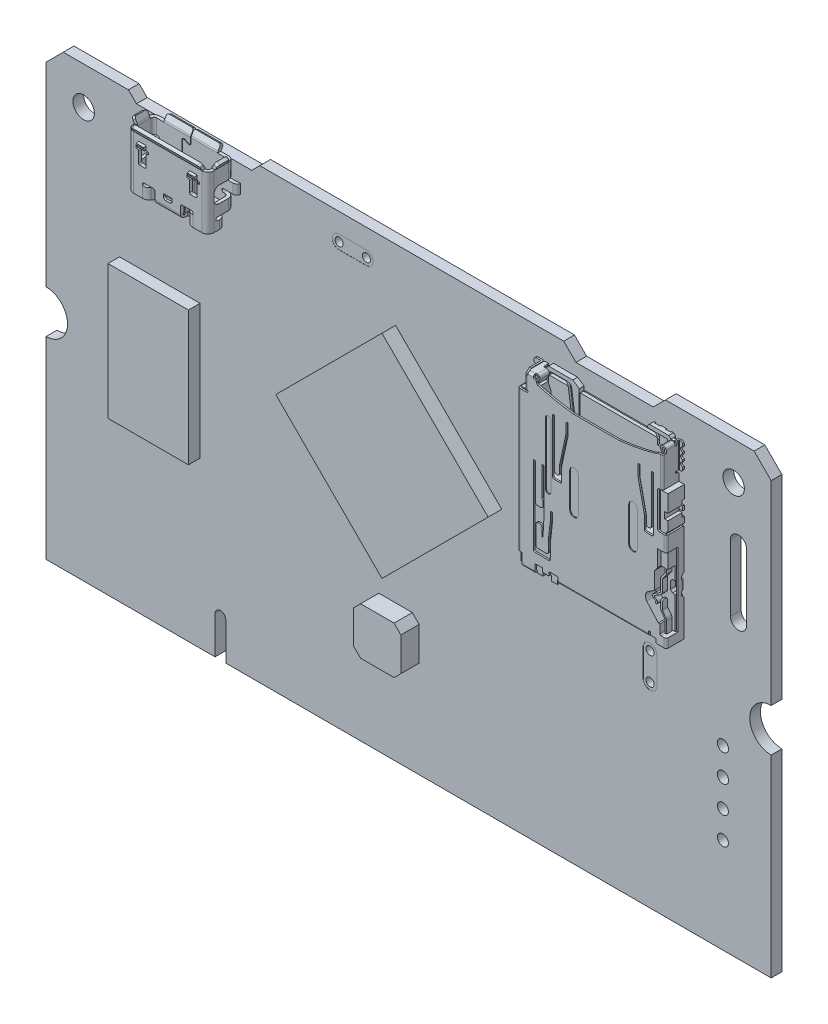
SolidWorks part; units mm, degrees
other "<475890001>-<Body-Move/Copy2>"
other "<microsd_card_slot>-<Imported1>"
ref_plane "Front" through (0, 0, 0) normal (0, 0, 1) x (1, 0, 0)
ref_plane "Top" through (0, 0, 0) normal (0, 1, 0) x (1, 0, 0)
ref_plane "Right" through (0, 0, 0) normal (1, 0, 0) x (0, 0, -1)
sketch "Sketch2" plane through (0, 0, 0) normal (0, 0, 1) x (1, 0, 0)
  line L0 (33.8, 0) -> (-17.05, 0)
  line L1 (-17.05, 0) -> (-17.05, 3.5)
  line L2 (-18.05, 3.5) -> (-18.05, 0)
  line L3 (-18.05, 0) -> (-33.8, 0)
  line L4 (-33.8, 0) -> (-33.8, 18)
  line L5 (-33.8, 22) -> (-33.8, 40.15)
  line L6 (-33.8, 40.15) -> (-32.2, 41.75)
  line L7 (-32.2, 41.75) -> (-26.125, 41.75)
  line L8 (-26.125, 41.75) -> (-25.375, 41)
  line L9 (-25.375, 41) -> (-14.625, 41)
  line L10 (-14.625, 41) -> (-13.875, 41.75)
  line L11 (-13.875, 41.75) -> (14.4595, 41.75)
  line L12 (14.4595, 41.75) -> (15.597, 40.6025)
  line L13 (15.597, 40.6025) -> (22.8, 40.6025)
  line L14 (22.8, 40.6025) -> (23.9475, 41.75)
  line L15 (23.9475, 41.75) -> (32.2078, 41.75)
  line L16 (32.2078, 41.75) -> (33.8, 40.1578)
  line L17 (33.8, 40.1578) -> (33.8, 22)
  line L18 (33.8, 18) -> (33.8, 0)
  line L19 (33.8, 0) -> (33.8, 18)
  line L20 (31.8, 20) -> (31.8, 14)
  line L21 (31.8, 14) -> (32.8, 14)
  line L22 (32.8, 14) -> (32.8, 0)
  line L23 (32.8, 0) -> (33.8, 0)
  line L24 (33.8, 0) -> (33.8, 18)
  line L25 (31.8, 20) -> (31.8, 14)
  line L26 (31.8, 14) -> (32.8, 14)
  line L27 (32.8, 14) -> (32.8, 0)
  line L28 (32.8, 0) -> (33.8, 0)
  line L29 (33.8, 0) -> (33.8, 18)
  line L30 (31.8, 20) -> (31.8, 14)
  line L31 (31.8, 14) -> (32.8, 14)
  line L32 (32.8, 14) -> (32.8, 0)
  line L33 (32.8, 0) -> (33.8, 0)
  line L34 (33.8, 0) -> (33.8, 18)
  line L35 (31.8, 20) -> (31.8, 14)
  line L36 (31.8, 14) -> (32.8, 14)
  line L37 (32.8, 14) -> (32.8, 0)
  line L38 (32.8, 0) -> (33.8, 0)
  line L39 (33.8, 0) -> (33.8, 18)
  line L40 (31.8, 20) -> (31.8, 14)
  line L41 (31.8, 14) -> (32.8, 14)
  line L42 (32.8, 14) -> (32.8, 0)
  line L43 (32.8, 0) -> (33.8, 0)
  line L44 (-33.8, 0) -> (-33.8, 18)
  line L45 (-31.8, 20) -> (-31.8, 14)
  line L46 (-31.8, 14) -> (-32.8, 14)
  line L47 (-32.8, 14) -> (-32.8, 0)
  line L48 (-32.8, 0) -> (-33.8, 0)
  line L49 (-33.8, 0) -> (-33.8, 18)
  line L50 (-31.8, 20) -> (-31.8, 14)
  line L51 (-31.8, 14) -> (-32.8, 14)
  line L52 (-32.8, 14) -> (-32.8, 0)
  line L53 (-32.8, 0) -> (-33.8, 0)
  line L54 (-33.8, 0) -> (-33.8, 18)
  line L55 (-31.8, 20) -> (-31.8, 14)
  line L56 (-31.8, 14) -> (-32.8, 14)
  line L57 (-32.8, 14) -> (-32.8, 0)
  line L58 (-32.8, 0) -> (-33.8, 0)
  line L59 (-33.8, 0) -> (-33.8, 18)
  line L60 (-31.8, 20) -> (-31.8, 14)
  line L61 (-31.8, 14) -> (-32.8, 14)
  line L62 (-32.8, 14) -> (-32.8, 0)
  line L63 (-32.8, 0) -> (-33.8, 0)
  line L64 (-33.8, 0) -> (-33.8, 18)
  line L65 (-31.8, 20) -> (-31.8, 14)
  line L66 (-31.8, 14) -> (-32.8, 14)
  line L67 (-32.8, 14) -> (-32.8, 0)
  line L68 (-32.8, 0) -> (-33.8, 0)
  line L69 (-30.8, 20) -> (-30.8, 4)
  line L70 (-30.8, 4) -> (-20, 4)
  line L71 (-20, 4) -> (-20, 4.2)
  line L72 (-20, 4.2) -> (-16, 4.2)
  line L73 (-16, 4.2) -> (-16, 4)
  line L74 (-16, 4) -> (0, 4)
  line L75 (0, 4) -> (0, 0)
  line L76 (0, 0) -> (-32.8, 0)
  line L77 (-32.8, 0) -> (-32.8, 14)
  line L78 (-32.8, 14) -> (-31.8, 14)
  line L79 (-31.8, 14) -> (-31.8, 20)
  line L80 (-33.8, 22) -> (-33.8, 31.75)
  line L81 (-33.8, 31.75) -> (-31.8, 31.75)
  line L82 (-31.8, 31.75) -> (-31.8, 22.2362)
  line L83 (-30.8, 20) -> (-30.8, 4)
  line L84 (-30.8, 4) -> (-20, 4)
  line L85 (-20, 4) -> (-20, 4.2)
  line L86 (-20, 4.2) -> (-16, 4.2)
  line L87 (-16, 4.2) -> (-16, 4)
  line L88 (-16, 4) -> (0, 4)
  line L89 (0, 4) -> (0, 0)
  line L90 (0, 0) -> (-32.8, 0)
  line L91 (-32.8, 0) -> (-32.8, 14)
  line L92 (-32.8, 14) -> (-31.8, 14)
  line L93 (-31.8, 14) -> (-31.8, 20)
  line L94 (-33.8, 22) -> (-33.8, 31.75)
  line L95 (-33.8, 31.75) -> (-31.8, 31.75)
  line L96 (-31.8, 31.75) -> (-31.8, 22.2362)
  line L97 (-30.8, 20) -> (-30.8, 4)
  line L98 (-30.8, 4) -> (-20, 4)
  line L99 (-20, 4) -> (-20, 4.2)
  line L100 (-20, 4.2) -> (-16, 4.2)
  line L101 (-16, 4.2) -> (-16, 4)
  line L102 (-16, 4) -> (0, 4)
  line L103 (0, 4) -> (0, 0)
  line L104 (0, 0) -> (-32.8, 0)
  line L105 (-32.8, 0) -> (-32.8, 14)
  line L106 (-32.8, 14) -> (-31.8, 14)
  line L107 (-31.8, 14) -> (-31.8, 20)
  line L108 (-33.8, 22) -> (-33.8, 31.75)
  line L109 (-33.8, 31.75) -> (-31.8, 31.75)
  line L110 (-31.8, 31.75) -> (-31.8, 22.2362)
  line L111 (30.8, 20) -> (30.8, 4)
  line L112 (30.8, 4) -> (0, 4)
  line L113 (0, 4) -> (0, 0)
  line L114 (0, 0) -> (32.8, 0)
  line L115 (32.8, 0) -> (32.8, 14)
  line L116 (32.8, 14) -> (31.8, 14)
  line L117 (31.8, 14) -> (31.8, 20)
  line L118 (33.8, 22) -> (33.8, 31.75)
  line L119 (33.8, 31.75) -> (31.8, 31.75)
  line L120 (31.8, 31.75) -> (31.8, 22.2362)
  line L121 (30.8, 20) -> (30.8, 4)
  line L122 (30.8, 4) -> (0, 4)
  line L123 (0, 4) -> (0, 0)
  line L124 (0, 0) -> (32.8, 0)
  line L125 (32.8, 0) -> (32.8, 14)
  line L126 (32.8, 14) -> (31.8, 14)
  line L127 (31.8, 14) -> (31.8, 20)
  line L128 (33.8, 22) -> (33.8, 31.75)
  line L129 (33.8, 31.75) -> (31.8, 31.75)
  line L130 (31.8, 31.75) -> (31.8, 22.2362)
  line L131 (30.8, 20) -> (30.8, 4)
  line L132 (30.8, 4) -> (0, 4)
  line L133 (0, 4) -> (0, 0)
  line L134 (0, 0) -> (32.8, 0)
  line L135 (32.8, 0) -> (32.8, 14)
  line L136 (32.8, 14) -> (31.8, 14)
  line L137 (31.8, 14) -> (31.8, 20)
  line L138 (33.8, 22) -> (33.8, 31.75)
  line L139 (33.8, 31.75) -> (31.8, 31.75)
  line L140 (31.8, 31.75) -> (31.8, 22.2362)
  line L141 (-24.93, 41.47) -> (-24.93, 37.77)
  line L142 (-24.93, 37.77) -> (-22.78, 35.62)
  line L143 (-22.78, 35.62) -> (-17.43, 35.62)
  line L144 (-17.43, 35.62) -> (-15.055, 37.995)
  line L145 (-15.055, 37.995) -> (-15.055, 41.47)
  line L146 (-15.055, 41.47) -> (-24.93, 41.47)
  line L147 (33.8, 0) -> (33.8007, 0)
  line L148 (32.2078, 41.75) -> (32.2085, 41.75)
  line L149 (-33.8, 40.15) -> (-33.7993, 40.15)
  line L150 (33.8, 40.1578) -> (33.8007, 40.1578)
  line L151 (33.8, 0) -> (33.8007, 0)
  line L152 (32.2078, 41.75) -> (32.2085, 41.75)
  line L153 (-33.8, 40.15) -> (-33.7993, 40.15)
  line L154 (33.8, 40.1578) -> (33.8007, 40.1578)
  line L155 (8.6, 34.5) -> (9, 34.5)
  line L156 (9, 34.5) -> (9, 37.5)
  line L157 (9, 37.5) -> (8.6, 37.5)
  line L158 (8.6, 37.5) -> (8.6, 34.5)
  line L159 (7.125, 36.65) -> (8.175, 36.65)
  line L160 (8.175, 36.65) -> (8.175, 37.25)
  line L161 (8.175, 37.25) -> (7.125, 37.25)
  line L162 (7.125, 37.25) -> (7.125, 36.65)
  line L163 (7.125, 34.75) -> (8.175, 34.75)
  line L164 (8.175, 34.75) -> (8.175, 35.35)
  line L165 (8.175, 35.35) -> (7.125, 35.35)
  line L166 (7.125, 35.35) -> (7.125, 34.75)
  line L167 (9.425, 35.7) -> (10.475, 35.7)
  line L168 (10.475, 35.7) -> (10.475, 36.3)
  line L169 (10.475, 36.3) -> (9.425, 36.3)
  line L170 (9.425, 36.3) -> (9.425, 35.7)
  line L171 (-3.9477, 38.6503) -> (-6.4877, 38.6503)
  line L172 (-6.4877, 39.9203) -> (-3.9477, 39.9203)
  line L173 (-3.9477, 38.3709) -> (-6.4877, 38.3709)
  line L174 (-6.4877, 40.1997) -> (-3.9477, 40.1997)
  line L175 (21.865, 18.23) -> (21.865, 20.77)
  line L176 (23.135, 20.77) -> (23.135, 18.23)
  line L177 (21.5856, 18.23) -> (21.5856, 20.77)
  line L178 (23.4144, 20.77) -> (23.4144, 18.23)
  line L179 (8.34, 40.55) -> (9.27, 40.55)
  line L180 (8.55, 41.55) -> (9.05, 41.55)
  line L181 (8.25, 40.3) -> (8.25, 41.3)
  line L182 (8.25, 41.3) -> (7.5, 41.3)
  line L183 (7.5, 41.3) -> (7.5, 40.3)
  line L184 (7.5, 40.3) -> (8.25, 40.3)
  line L185 (10.1, 40.3) -> (10.1, 41.3)
  line L186 (10.1, 41.3) -> (9.35, 41.3)
  line L187 (9.35, 41.3) -> (9.35, 40.3)
  line L188 (9.35, 40.3) -> (10.1, 40.3)
  line L189 (12.0759, 18.3556) -> (13.3134, 17.1182)
  line L190 (13.3134, 17.1182) -> (14.7276, 18.5324)
  line L191 (14.7276, 18.5324) -> (13.4902, 19.7699)
  line L192 (13.4902, 19.7699) -> (12.0759, 18.3556)
  line L193 (11.9345, 18.5678) -> (13.278, 19.9113)
  line L194 (13.278, 19.9113) -> (12.5002, 20.6891)
  line L195 (12.5002, 20.6891) -> (11.1567, 19.3456)
  line L196 (11.1567, 19.3456) -> (11.9345, 18.5678)
  line L197 (14.3387, 16.1636) -> (15.6822, 17.5071)
  line L198 (15.6822, 17.5071) -> (14.9044, 18.2849)
  line L199 (14.9044, 18.2849) -> (13.5609, 16.9414)
  line L200 (13.5609, 16.9414) -> (14.3387, 16.1636)
  line L201 (24.95, 35.7) -> (14.8, 35.7)
  line L202 (14.8, 35.7) -> (14.8, 33.35)
  line L203 (14.8, 33.35) -> (15.15, 33.35)
  line L204 (15.15, 33.35) -> (15.15, 27.35)
  line L205 (15.15, 27.35) -> (20.8, 27.35)
  line L206 (20.8, 27.35) -> (20.8, 24.85)
  line L207 (20.8, 24.85) -> (23.85, 24.85)
  line L208 (23.85, 24.85) -> (23.85, 23.6)
  line L209 (23.85, 23.6) -> (25.95, 23.6)
  line L210 (25.95, 23.6) -> (25.95, 31.8)
  line L211 (25.95, 31.8) -> (24.7, 31.8)
  line L212 (24.7, 31.8) -> (24.7, 32.9)
  line L213 (24.7, 32.9) -> (25.95, 32.9)
  line L214 (25.95, 32.9) -> (25.95, 36.7)
  line L215 (25.95, 36.7) -> (24.95, 36.7)
  line L216 (24.95, 36.7) -> (24.95, 35.7)
  line L217 (24.95, 35.7) -> (14.8, 35.7)
  line L218 (14.8, 35.7) -> (14.8, 33.35)
  line L219 (14.8, 33.35) -> (15.15, 33.35)
  line L220 (15.15, 33.35) -> (15.15, 27.35)
  line L221 (15.15, 27.35) -> (20.8, 27.35)
  line L222 (20.8, 27.35) -> (20.8, 24.85)
  line L223 (20.8, 24.85) -> (23.85, 24.85)
  line L224 (23.85, 24.85) -> (23.85, 23.6)
  line L225 (23.85, 23.6) -> (25.95, 23.6)
  line L226 (25.95, 23.6) -> (25.95, 31.8)
  line L227 (25.95, 31.8) -> (24.7, 31.8)
  line L228 (24.7, 31.8) -> (24.7, 32.9)
  line L229 (24.7, 32.9) -> (25.95, 32.9)
  line L230 (25.95, 32.9) -> (25.95, 36.7)
  line L231 (25.95, 36.7) -> (24.95, 36.7)
  line L232 (24.95, 36.7) -> (24.95, 35.7)
  line L233 (24.95, 35.7) -> (14.8, 35.7)
  line L234 (14.8, 35.7) -> (14.8, 33.35)
  line L235 (14.8, 33.35) -> (15.15, 33.35)
  line L236 (15.15, 33.35) -> (15.15, 27.35)
  line L237 (15.15, 27.35) -> (20.8, 27.35)
  line L238 (20.8, 27.35) -> (20.8, 24.85)
  line L239 (20.8, 24.85) -> (23.85, 24.85)
  line L240 (23.85, 24.85) -> (23.85, 23.6)
  line L241 (23.85, 23.6) -> (25.95, 23.6)
  line L242 (25.95, 23.6) -> (25.95, 31.8)
  line L243 (25.95, 31.8) -> (24.7, 31.8)
  line L244 (24.7, 31.8) -> (24.7, 32.9)
  line L245 (24.7, 32.9) -> (25.95, 32.9)
  line L246 (25.95, 32.9) -> (25.95, 36.7)
  line L247 (25.95, 36.7) -> (24.95, 36.7)
  line L248 (24.95, 36.7) -> (24.95, 35.7)
  line L249 (24.95, 35.7) -> (14.8, 35.7)
  line L250 (14.8, 35.7) -> (14.8, 33.35)
  line L251 (14.8, 33.35) -> (15.15, 33.35)
  line L252 (15.15, 33.35) -> (15.15, 27.35)
  line L253 (15.15, 27.35) -> (20.8, 27.35)
  line L254 (20.8, 27.35) -> (20.8, 24.85)
  line L255 (20.8, 24.85) -> (23.85, 24.85)
  line L256 (23.85, 24.85) -> (23.85, 23.6)
  line L257 (23.85, 23.6) -> (25.95, 23.6)
  line L258 (25.95, 23.6) -> (25.95, 31.8)
  line L259 (25.95, 31.8) -> (24.7, 31.8)
  line L260 (24.7, 31.8) -> (24.7, 32.9)
  line L261 (24.7, 32.9) -> (25.95, 32.9)
  line L262 (25.95, 32.9) -> (25.95, 36.7)
  line L263 (25.95, 36.7) -> (24.95, 36.7)
  line L264 (24.95, 36.7) -> (24.95, 35.7)
  line L265 (12.4, 35.2) -> (11.55, 35.2)
  line L266 (11.55, 35.2) -> (11.55, 37.15)
  line L267 (11.55, 37.15) -> (12.4, 37.15)
  line L268 (12.4, 37.15) -> (12.4, 35.2)
  line L269 (12.4, 35.2) -> (11.55, 35.2)
  line L270 (11.55, 35.2) -> (11.55, 37.15)
  line L271 (11.55, 37.15) -> (12.4, 37.15)
  line L272 (12.4, 37.15) -> (12.4, 35.2)
  line L273 (12.4, 35.2) -> (11.55, 35.2)
  line L274 (11.55, 35.2) -> (11.55, 37.15)
  line L275 (11.55, 37.15) -> (12.4, 37.15)
  line L276 (12.4, 37.15) -> (12.4, 35.2)
  line L277 (12.4, 35.2) -> (11.55, 35.2)
  line L278 (11.55, 35.2) -> (11.55, 37.15)
  line L279 (11.55, 37.15) -> (12.4, 37.15)
  line L280 (12.4, 37.15) -> (12.4, 35.2)
  line L281 (25.6, 39.775) -> (11.9, 39.775)
  line L282 (11.9, 23.3) -> (11.9, 37.4)
  line L283 (25.6, 33.15) -> (25.6, 37.25)
  line L284 (25.6, 23.3) -> (25.6, 31.55)
  line L285 (25.6, 23.3) -> (11.9, 23.3)
  line L286 (25.851, 37.5) -> (24.601, 37.5)
  line L287 (24.501, 37.6) -> (24.501, 38.8)
  line L288 (24.601, 38.9) -> (25.851, 38.9)
  line L289 (25.951, 38.8) -> (25.951, 37.6)
  line L290 (12.65, 39.2) -> (12.65, 37.8)
  line L291 (12.55, 37.7) -> (11.65, 37.7)
  line L292 (11.55, 37.8) -> (11.55, 39.2)
  line L293 (11.65, 39.3) -> (12.55, 39.3)
  line L294 (25.85, 31.9) -> (24.9, 31.9)
  line L295 (24.8, 32) -> (24.8, 32.7)
  line L296 (24.9, 32.8) -> (25.85, 32.8)
  line L297 (25.95, 32.7) -> (25.95, 32)
  line L298 (-19.375, 34.8) -> (-19.975, 34.8)
  line L299 (-18.075, 34.8) -> (-17.875, 34.8)
  line L300 (-17.875, 34.8) -> (-17.875, 32)
  line L301 (-17.875, 32) -> (-18.975, 32)
  line L302 (-21.275, 34.8) -> (-21.475, 34.8)
  line L303 (-21.475, 34.8) -> (-21.475, 32)
  line L304 (-21.475, 32) -> (-20.375, 32)
  line L305 (-19.17, 35.1) -> (-19.17, 33.7)
  line L306 (-19.17, 33.7) -> (-18.27, 33.7)
  line L307 (-18.27, 33.7) -> (-18.27, 35.1)
  line L308 (-18.27, 35.1) -> (-19.17, 35.1)
  line L309 (-21.08, 35.1) -> (-21.08, 33.7)
  line L310 (-21.08, 33.7) -> (-20.18, 33.7)
  line L311 (-20.18, 33.7) -> (-20.18, 35.1)
  line L312 (-20.18, 35.1) -> (-21.08, 35.1)
  line L313 (-20.125, 33.1) -> (-20.125, 31.7)
  line L314 (-20.125, 31.7) -> (-19.225, 31.7)
  line L315 (-19.225, 31.7) -> (-19.225, 33.1)
  line L316 (-19.225, 33.1) -> (-20.125, 33.1)
  line L317 (-24.1, 38.3) -> (-24.1, 35.8)
  line L318 (-24.1, 35.8) -> (-22.9, 35.8)
  line L319 (-18.9, 37.475) -> (-18.9, 36.125)
  line L320 (-18.9, 36.125) -> (-18.5, 36.125)
  line L321 (-18.5, 36.125) -> (-18.5, 37.475)
  line L322 (-18.5, 37.475) -> (-18.9, 37.475)
  line L323 (-19.55, 37.475) -> (-19.55, 36.125)
  line L324 (-19.55, 36.125) -> (-19.15, 36.125)
  line L325 (-19.15, 36.125) -> (-19.15, 37.475)
  line L326 (-19.15, 37.475) -> (-19.55, 37.475)
  line L327 (-20.2, 37.475) -> (-20.2, 36.125)
  line L328 (-20.2, 36.125) -> (-19.8, 36.125)
  line L329 (-19.8, 36.125) -> (-19.8, 37.475)
  line L330 (-19.8, 37.475) -> (-20.2, 37.475)
  line L331 (-20.85, 37.475) -> (-20.85, 36.125)
  line L332 (-20.85, 36.125) -> (-20.45, 36.125)
  line L333 (-20.45, 36.125) -> (-20.45, 37.475)
  line L334 (-20.45, 37.475) -> (-20.85, 37.475)
  line L335 (-21.5, 37.475) -> (-21.5, 36.125)
  line L336 (-21.5, 36.125) -> (-21.1, 36.125)
  line L337 (-21.1, 36.125) -> (-21.1, 37.475)
  line L338 (-21.1, 37.475) -> (-21.5, 37.475)
  line L339 (-18.35, 36.525) -> (-18.35, 36.425)
  line L340 (-18.35, 36.425) -> (-17.2, 36.425)
  line L341 (-17.2, 36.425) -> (-17.2, 36.525)
  line L342 (-17.2, 36.525) -> (-18.35, 36.525)
  line L343 (-22.8, 36.525) -> (-22.8, 36.425)
  line L344 (-22.8, 36.425) -> (-21.65, 36.425)
  line L345 (-21.65, 36.425) -> (-21.65, 36.525)
  line L346 (-21.65, 36.525) -> (-22.8, 36.525)
  line L347 (-19.75, 40.425) -> (-19.75, 38.525)
  line L348 (-19.75, 38.525) -> (-17.95, 38.525)
  line L349 (-17.95, 38.525) -> (-17.95, 40.425)
  line L350 (-17.95, 40.425) -> (-19.75, 40.425)
  line L351 (-22.05, 40.425) -> (-22.05, 38.525)
  line L352 (-22.05, 38.525) -> (-20.25, 38.525)
  line L353 (-20.25, 38.525) -> (-20.25, 40.425)
  line L354 (-20.25, 40.425) -> (-22.05, 40.425)
  line L355 (-16.51, 39.825) -> (-16.51, 39.125)
  line L356 (-16.51, 39.125) -> (-15.31, 39.125)
  line L357 (-15.31, 39.125) -> (-15.31, 39.825)
  line L358 (-15.31, 39.825) -> (-16.51, 39.825)
  line L359 (-15.91, 38.525) -> (-17.4, 38.525)
  line L360 (-17.4, 38.525) -> (-17.4, 40.425)
  line L361 (-17.4, 40.425) -> (-15.91, 40.425)
  line L362 (-15.91, 40.425) -> (-15.91, 38.525)
  line L363 (-24.69, 39.825) -> (-24.69, 39.125)
  line L364 (-24.69, 39.125) -> (-23.49, 39.125)
  line L365 (-23.49, 39.125) -> (-23.49, 39.825)
  line L366 (-23.49, 39.825) -> (-24.69, 39.825)
  line L367 (-24.09, 40.425) -> (-22.6, 40.425)
  line L368 (-22.6, 40.425) -> (-22.6, 38.525)
  line L369 (-22.6, 38.525) -> (-24.09, 38.525)
  line L370 (-24.09, 38.525) -> (-24.09, 40.425)
  line L371 (-19.45, 27.85) -> (-26.95, 27.85)
  line L372 (-26.95, 27.85) -> (-26.95, 15.35)
  line L373 (-26.95, 15.35) -> (-19.45, 15.35)
  line L374 (-19.45, 15.35) -> (-19.45, 27.85)
  line L375 (-1.2177, 35.1848) -> (8.6818, 25.2853)
  line L376 (8.6818, 25.2853) -> (-1.2177, 15.3858)
  line L377 (-1.2177, 15.3858) -> (-11.1172, 25.2853)
  line L378 (-11.1172, 25.2853) -> (-1.2177, 35.1848)
  line L379 (-24.95, 33.7) -> (-24.95, 33.1)
  line L380 (-24.95, 33.1) -> (-22.05, 33.1)
  line L381 (-22.05, 33.1) -> (-22.05, 33.7)
  line L382 (-22.05, 33.7) -> (-24.95, 33.7)
  line L383 (-22.875, 35.075) -> (-22.875, 34.025)
  line L384 (-22.875, 34.025) -> (-22.225, 34.025)
  line L385 (-22.225, 34.025) -> (-22.225, 35.075)
  line L386 (-22.225, 35.075) -> (-22.875, 35.075)
  line L387 (-24.775, 35.075) -> (-24.775, 34.025)
  line L388 (-24.775, 34.025) -> (-24.125, 34.025)
  line L389 (-24.125, 34.025) -> (-24.125, 35.075)
  line L390 (-24.125, 35.075) -> (-24.775, 35.075)
  line L391 (-23.825, 32.775) -> (-23.825, 31.725)
  line L392 (-23.825, 31.725) -> (-23.175, 31.725)
  line L393 (-23.175, 31.725) -> (-23.175, 32.775)
  line L394 (-23.175, 32.775) -> (-23.825, 32.775)
  line L395 (13.1366, 14.0423) -> (12.7123, 13.618)
  line L396 (9.6011, 17.5778) -> (9.1768, 17.1536)
  line L397 (11.6517, 17.3657) -> (12.9245, 16.0929)
  line L398 (9.3889, 15.1029) -> (10.6617, 13.8301)
  line L399 (12.5002, 15.1737) -> (13.6316, 14.0423)
  line L400 (13.6316, 14.0423) -> (14.5508, 14.9615)
  line L401 (14.5508, 14.9615) -> (13.4194, 16.0929)
  line L402 (13.4194, 16.0929) -> (12.5002, 15.1737)
  line L403 (9.6011, 18.0728) -> (10.7324, 16.9414)
  line L404 (10.7324, 16.9414) -> (11.6517, 17.8607)
  line L405 (11.6517, 17.8607) -> (10.5203, 18.992)
  line L406 (10.5203, 18.992) -> (9.6011, 18.0728)
  line L407 (7.7626, 16.2343) -> (8.894, 15.1029)
  line L408 (8.894, 15.1029) -> (9.8132, 16.0222)
  line L409 (9.8132, 16.0222) -> (8.6818, 17.1536)
  line L410 (8.6818, 17.1536) -> (7.7626, 16.2343)
  line L411 (10.6617, 13.3352) -> (11.7931, 12.2038)
  line L412 (11.7931, 12.2038) -> (12.7123, 13.123)
  line L413 (12.7123, 13.123) -> (11.581, 14.2544)
  line L414 (11.581, 14.2544) -> (10.6617, 13.3352)
  line L415 (-11.5061, 17.1182) -> (-10.7282, 16.3404)
  line L416 (-10.7282, 16.3404) -> (-10.5161, 16.5525)
  line L417 (-10.5161, 16.5525) -> (-11.2939, 17.3303)
  line L418 (-11.2939, 17.3303) -> (-11.5061, 17.1182)
  line L419 (-10.7282, 16.3404) -> (-10.5161, 16.5525)
  line L420 (-11.6475, 17.6839) -> (-11.7182, 17.6132)
  line L421 (-11.7182, 17.6132) -> (-11.5768, 17.4718)
  line L422 (-11.5768, 17.4718) -> (-11.5061, 17.1182)
  line L423 (-11.5061, 17.1182) -> (-10.7282, 16.3404)
  line L424 (-11.6828, 17.6485) -> (-11.5768, 17.5425)
  line L425 (-11.5768, 17.5425) -> (-12.1425, 16.9768)
  line L426 (-12.1425, 16.9768) -> (-12.2485, 17.0828)
  line L427 (-12.2485, 17.0828) -> (-11.6828, 17.6485)
  line L428 (-11.9303, 16.6939) -> (-11.1525, 15.9161)
  line L429 (-11.1525, 15.9161) -> (-10.9404, 16.1283)
  line L430 (-10.9404, 16.1283) -> (-11.7182, 16.9061)
  line L431 (-11.7182, 16.9061) -> (-11.9303, 16.6939)
  line L432 (-10.9404, 16.1283) -> (-11.1525, 15.9161)
  line L433 (-12.2839, 17.0475) -> (-12.2132, 17.1182)
  line L434 (-12.2132, 17.1182) -> (-12.0717, 16.9768)
  line L435 (-12.0717, 16.9768) -> (-11.7182, 16.9061)
  line L436 (-11.7182, 16.9061) -> (-10.9404, 16.1283)
  line L437 (-29, 5) -> (-29, 5.5)
  line L438 (-30, 6) -> (-29.5, 6)
  line L439 (-29, 6.5) -> (-29, 7)
  line L440 (-28.5, 6) -> (-28, 6)
  line L441 (-28.6465, 6.3536) -> (-28.2929, 6.7071)
  line L442 (-29.321, 6.321) -> (-29.7071, 6.7071)
  line L443 (-29.7071, 5.2929) -> (-29.3535, 5.6464)
  line L444 (-28.2929, 5.2929) -> (-28.6465, 5.6464)
  line L445 (-32, 32) -> (-32, 32.5)
  line L446 (-33, 33) -> (-32.5, 33)
  line L447 (-32, 33.5) -> (-32, 34)
  line L448 (-31.5, 33) -> (-31, 33)
  line L449 (-31.6464, 33.3536) -> (-31.2929, 33.7071)
  line L450 (-32.321, 33.321) -> (-32.7071, 33.7071)
  line L451 (-32.7071, 32.2929) -> (-32.3535, 32.6465)
  line L452 (-31.2929, 32.2929) -> (-31.6464, 32.6465)
  line L453 (29.7071, 5.2929) -> (29.3535, 5.6464)
  line L454 (28.2929, 5.2929) -> (28.6465, 5.6464)
  line L455 (28.6465, 6.3536) -> (28.2929, 6.7071)
  line L456 (29.3535, 6.3536) -> (29.7071, 6.7071)
  line L457 (29, 6.5) -> (29, 7)
  line L458 (28.5461, 6) -> (28, 6)
  line L459 (29, 5) -> (29, 5.5)
  line L460 (30, 6) -> (29.5, 6)
  line L461 (1.1823, 8.1775) -> (-3.6177, 8.1775)
  line L462 (-3.6177, 8.1775) -> (-3.6177, 12.9775)
  line L463 (-3.6177, 12.9775) -> (1.1823, 12.9775)
  line L464 (1.1823, 12.9775) -> (1.1823, 8.1775)
  line L465 (0.2823, 12.1395) -> (0.2823, 9.0155)
  line L466 (0.2823, 9.0155) -> (0.9823, 9.0155)
  line L467 (0.9823, 9.0155) -> (0.9823, 12.1395)
  line L468 (0.9823, 12.1395) -> (0.2823, 12.1395)
  line L469 (0.9823, 11.7275) -> (0.2823, 11.7275)
  line L470 (0.2823, 11.7275) -> (-0.0677, 12.0775)
  line L471 (-0.0677, 12.0775) -> (-0.4677, 12.0775)
  line L472 (-0.4677, 12.0775) -> (-0.4677, 12.7775)
  line L473 (-0.4677, 12.7775) -> (0.3443, 12.7775)
  line L474 (0.3443, 12.7775) -> (0.9823, 12.1395)
  line L475 (0.9823, 12.1395) -> (0.9823, 11.7275)
  line L476 (0.9823, 9.4275) -> (0.2823, 9.4275)
  line L477 (0.2823, 9.4275) -> (-0.0677, 9.0775)
  line L478 (-0.0677, 9.0775) -> (-0.4677, 9.0775)
  line L479 (-0.4677, 9.0775) -> (-0.4677, 8.3775)
  line L480 (-0.4677, 8.3775) -> (0.3443, 8.3775)
  line L481 (0.3443, 8.3775) -> (0.9823, 9.0155)
  line L482 (0.9823, 9.0155) -> (0.9823, 9.4275)
  line L483 (-3.4177, 12.1395) -> (-3.4177, 9.0155)
  line L484 (-3.4177, 9.0155) -> (-2.7177, 9.0155)
  line L485 (-2.7177, 9.0155) -> (-2.7177, 12.1395)
  line L486 (-2.7177, 12.1395) -> (-3.4177, 12.1395)
  line L487 (-3.4177, 9.4275) -> (-2.7177, 9.4275)
  line L488 (-2.7177, 9.4275) -> (-2.3677, 9.0775)
  line L489 (-2.3677, 9.0775) -> (-1.9677, 9.0775)
  line L490 (-1.9677, 9.0775) -> (-1.9677, 8.3775)
  line L491 (-1.9677, 8.3775) -> (-2.7797, 8.3775)
  line L492 (-2.7797, 8.3775) -> (-3.4177, 9.0155)
  line L493 (-3.4177, 9.0155) -> (-3.4177, 9.4275)
  line L494 (-3.4177, 11.7275) -> (-2.7177, 11.7275)
  line L495 (-2.7177, 11.7275) -> (-2.3677, 12.0775)
  line L496 (-2.3677, 12.0775) -> (-1.9677, 12.0775)
  line L497 (-1.9677, 12.0775) -> (-1.9677, 12.7775)
  line L498 (-1.9677, 12.7775) -> (-2.7797, 12.7775)
  line L499 (-2.7797, 12.7775) -> (-3.4177, 12.1395)
  line L500 (-3.4177, 12.1395) -> (-3.4177, 11.7275)
  line L501 (1.9184, 16.6409) -> (3.1487, 15.4105)
  line L502 (3.1487, 15.4105) -> (3.5518, 15.8136)
  line L503 (3.5518, 15.8136) -> (2.3214, 17.0439)
  line L504 (2.3214, 17.0439) -> (1.9184, 16.6409)
  line L505 (1.3668, 16.0894) -> (2.5972, 14.859)
  line L506 (2.5972, 14.859) -> (3.0002, 15.262)
  line L507 (3.0002, 15.262) -> (1.7699, 16.4924)
  line L508 (1.7699, 16.4924) -> (1.3668, 16.0894)
  line L509 (1.586, 13.8478) -> (0.3557, 15.0782)
  line L510 (0.3557, 15.0782) -> (-0.0474, 14.6752)
  line L511 (-0.0474, 14.6752) -> (1.183, 13.4448)
  line L512 (1.183, 13.4448) -> (1.586, 13.8478)
  line L513 (2.1376, 14.3994) -> (0.9072, 15.6297)
  line L514 (0.9072, 15.6297) -> (0.5041, 15.2267)
  line L515 (0.5041, 15.2267) -> (1.7345, 13.9963)
  line L516 (1.7345, 13.9963) -> (2.1376, 14.3994)
  line L517 (2.3543, 6.1012) -> (2.3543, 7.8412)
  line L518 (2.3543, 7.8412) -> (1.7843, 7.8412)
  line L519 (1.7843, 7.8412) -> (1.7843, 6.1012)
  line L520 (1.7843, 6.1012) -> (2.3543, 6.1012)
  line L521 (3.1343, 6.1012) -> (3.1343, 7.8412)
  line L522 (3.1343, 7.8412) -> (2.5643, 7.8412)
  line L523 (2.5643, 7.8412) -> (2.5643, 6.1012)
  line L524 (2.5643, 6.1012) -> (3.1343, 6.1012)
  line L525 (-22.33, 13.095) -> (-24.07, 13.095)
  line L526 (-24.07, 13.095) -> (-24.07, 12.525)
  line L527 (-24.07, 12.525) -> (-22.33, 12.525)
  line L528 (-22.33, 12.525) -> (-22.33, 13.095)
  line L529 (-22.33, 13.875) -> (-24.07, 13.875)
  line L530 (-24.07, 13.875) -> (-24.07, 13.305)
  line L531 (-24.07, 13.305) -> (-22.33, 13.305)
  line L532 (-22.33, 13.305) -> (-22.33, 13.875)
  line L533 (-22.33, 10.995) -> (-24.07, 10.995)
  line L534 (-24.07, 10.995) -> (-24.07, 10.425)
  line L535 (-24.07, 10.425) -> (-22.33, 10.425)
  line L536 (-22.33, 10.425) -> (-22.33, 10.995)
  line L537 (-22.33, 11.775) -> (-24.07, 11.775)
  line L538 (-24.07, 11.775) -> (-24.07, 11.205)
  line L539 (-24.07, 11.205) -> (-22.33, 11.205)
  line L540 (-22.33, 11.205) -> (-22.33, 11.775)
  line L541 (3.2414, 17.9747) -> (4.4718, 16.7444)
  line L542 (4.4718, 16.7444) -> (4.8748, 17.1474)
  line L543 (4.8748, 17.1474) -> (3.6444, 18.3778)
  line L544 (3.6444, 18.3778) -> (3.2414, 17.9747)
  line L545 (2.6899, 17.4232) -> (3.9202, 16.1928)
  line L546 (3.9202, 16.1928) -> (4.3233, 16.5958)
  line L547 (4.3233, 16.5958) -> (3.0929, 17.8262)
  line L548 (3.0929, 17.8262) -> (2.6899, 17.4232)
  line L549 (6.37, 36.895) -> (4.63, 36.895)
  line L550 (4.63, 36.895) -> (4.63, 36.325)
  line L551 (4.63, 36.325) -> (6.37, 36.325)
  line L552 (6.37, 36.325) -> (6.37, 36.895)
  line L553 (6.37, 37.675) -> (4.63, 37.675)
  line L554 (4.63, 37.675) -> (4.63, 37.105)
  line L555 (4.63, 37.105) -> (6.37, 37.105)
  line L556 (6.37, 37.105) -> (6.37, 37.675)
  line L557 (-8.0306, 18.939) -> (-9.261, 20.1694)
  line L558 (-9.261, 20.1694) -> (-9.664, 19.7663)
  line L559 (-9.664, 19.7663) -> (-8.4337, 18.5359)
  line L560 (-8.4337, 18.5359) -> (-8.0306, 18.939)
  line L561 (-7.4791, 19.4905) -> (-8.7095, 20.7209)
  line L562 (-8.7095, 20.7209) -> (-9.1125, 20.3179)
  line L563 (-9.1125, 20.3179) -> (-7.8821, 19.0875)
  line L564 (-7.8821, 19.0875) -> (-7.4791, 19.4905)
  line L565 (-4.9996, 6.1012) -> (-4.9996, 7.8412)
  line L566 (-4.9996, 7.8412) -> (-5.5696, 7.8412)
  line L567 (-5.5696, 7.8412) -> (-5.5696, 6.1012)
  line L568 (-5.5696, 6.1012) -> (-4.9996, 6.1012)
  line L569 (-4.2196, 6.1012) -> (-4.2196, 7.8412)
  line L570 (-4.2196, 7.8412) -> (-4.7896, 7.8412)
  line L571 (-4.7896, 7.8412) -> (-4.7896, 6.1012)
  line L572 (-4.7896, 6.1012) -> (-4.2196, 6.1012)
  line L573 (6.1727, 6.1012) -> (6.1727, 7.8412)
  line L574 (6.1727, 7.8412) -> (5.6027, 7.8412)
  line L575 (5.6027, 7.8412) -> (5.6027, 6.1012)
  line L576 (5.6027, 6.1012) -> (6.1727, 6.1012)
  line L577 (6.9527, 6.1012) -> (6.9527, 7.8412)
  line L578 (6.9527, 7.8412) -> (6.3827, 7.8412)
  line L579 (6.3827, 7.8412) -> (6.3827, 6.1012)
  line L580 (6.3827, 6.1012) -> (6.9527, 6.1012)
  line L581 (28.305, 25.87) -> (28.305, 24.13)
  line L582 (28.305, 24.13) -> (28.875, 24.13)
  line L583 (28.875, 24.13) -> (28.875, 25.87)
  line L584 (28.875, 25.87) -> (28.305, 25.87)
  line L585 (27.525, 25.87) -> (27.525, 24.13)
  line L586 (27.525, 24.13) -> (28.095, 24.13)
  line L587 (28.095, 24.13) -> (28.095, 25.87)
  line L588 (28.095, 25.87) -> (27.525, 25.87)
  line L589 (28.305, 23.37) -> (28.305, 21.63)
  line L590 (28.305, 21.63) -> (28.875, 21.63)
  line L591 (28.875, 21.63) -> (28.875, 23.37)
  line L592 (28.875, 23.37) -> (28.305, 23.37)
  line L593 (27.525, 23.37) -> (27.525, 21.63)
  line L594 (27.525, 21.63) -> (28.095, 21.63)
  line L595 (28.095, 21.63) -> (28.095, 23.37)
  line L596 (28.095, 23.37) -> (27.525, 23.37)
  line L597 (9.0814, 9.5345) -> (7.851, 10.7648)
  line L598 (7.851, 10.7648) -> (7.4479, 10.3618)
  line L599 (7.4479, 10.3618) -> (8.6783, 9.1314)
  line L600 (8.6783, 9.1314) -> (9.0814, 9.5345)
  line L601 (9.6329, 10.086) -> (8.4025, 11.3164)
  line L602 (8.4025, 11.3164) -> (7.9995, 10.9133)
  line L603 (7.9995, 10.9133) -> (9.2298, 9.683)
  line L604 (9.2298, 9.683) -> (9.6329, 10.086)
  line L605 (-33.8, 40.15) -> (-32.2, 41.75)
  line L606 (-32.2, 41.75) -> (-26.8, 41.75)
  line L607 (-26.8, 41.75) -> (-26.8, 38.25)
  line L608 (-30.3, 34.75) -> (-33.8, 34.75)
  line L609 (-33.8, 34.75) -> (-33.8, 40.15)
  line L610 (32.2, 41.75) -> (33.8, 40.15)
  line L611 (33.8, 40.15) -> (33.8, 34.75)
  line L612 (33.8, 34.75) -> (30.3, 34.75)
  line L613 (26.8, 38.25) -> (26.8, 41.75)
  line L614 (26.8, 41.75) -> (32.2, 41.75)
  line L615 (9.7071, 21.9265) -> (9.3536, 22.2801)
  line L616 (9.3536, 22.2801) -> (9.7071, 22.6336)
  line L617 (9.7071, 22.6336) -> (10.0607, 22.2801)
  line L618 (9.3925, 21.9301) -> (8.9894, 22.3331)
  line L619 (8.9894, 22.3331) -> (9.64, 22.9837)
  line L620 (9.64, 22.9837) -> (10.043, 22.5806)
  line L621 (10.043, 22.5806) -> (9.3925, 21.9301)
  line L622 (9.9723, 22.5099) -> (9.5693, 22.9129)
  line L623 (9.5693, 22.9129) -> (10.2198, 23.5635)
  line L624 (10.2198, 23.5635) -> (10.6228, 23.1604)
  line L625 (10.6228, 23.1604) -> (9.9723, 22.5099)
  line L626 (10.2764, 22.4887) -> (9.9228, 22.8422)
  line L627 (9.9228, 22.8422) -> (10.2764, 23.1958)
  line L628 (10.2764, 23.1958) -> (10.6299, 22.8422)
  line L629 (8.4379, 22.8847) -> (8.8409, 22.4816)
  line L630 (8.8409, 22.4816) -> (9.4915, 23.1321)
  line L631 (9.4915, 23.1321) -> (9.0884, 23.5352)
  line L632 (9.0884, 23.5352) -> (8.4379, 22.8847)
  line L633 (8.7914, 23.5493) -> (9.145, 23.1958)
  line L634 (9.145, 23.1958) -> (8.7914, 22.8422)
  line L635 (8.7914, 22.8422) -> (8.4379, 23.1958)
  line L636 (9.0177, 23.4645) -> (9.4208, 23.0614)
  line L637 (9.4208, 23.0614) -> (10.0713, 23.712)
  line L638 (10.0713, 23.712) -> (9.6683, 24.115)
  line L639 (9.6683, 24.115) -> (9.0177, 23.4645)
  line L640 (9.3571, 24.115) -> (9.7107, 23.7615)
  line L641 (9.7107, 23.7615) -> (9.3571, 23.4079)
  line L642 (9.3571, 23.4079) -> (9.0036, 23.7615)
  line L643 (6.8787, 19.0981) -> (6.5252, 19.4517)
  line L644 (6.5252, 19.4517) -> (6.8787, 19.8052)
  line L645 (6.8787, 19.8052) -> (7.2323, 19.4517)
  line L646 (6.564, 19.1016) -> (6.161, 19.5047)
  line L647 (6.161, 19.5047) -> (6.8115, 20.1552)
  line L648 (6.8115, 20.1552) -> (7.2146, 19.7522)
  line L649 (7.2146, 19.7522) -> (6.564, 19.1016)
  line L650 (7.1439, 19.6815) -> (6.7408, 20.0845)
  line L651 (6.7408, 20.0845) -> (7.3914, 20.7351)
  line L652 (7.3914, 20.7351) -> (7.7944, 20.332)
  line L653 (7.7944, 20.332) -> (7.1439, 19.6815)
  line L654 (7.4479, 19.6603) -> (7.0944, 20.0138)
  line L655 (7.0944, 20.0138) -> (7.4479, 20.3673)
  line L656 (7.4479, 20.3673) -> (7.8015, 20.0138)
  line L657 (5.6095, 20.0562) -> (6.0125, 19.6532)
  line L658 (6.0125, 19.6532) -> (6.6631, 20.3037)
  line L659 (6.6631, 20.3037) -> (6.26, 20.7068)
  line L660 (6.26, 20.7068) -> (5.6095, 20.0562)
  line L661 (5.963, 20.7209) -> (6.3166, 20.3673)
  line L662 (6.3166, 20.3673) -> (5.963, 20.0138)
  line L663 (5.963, 20.0138) -> (5.6095, 20.3673)
  line L664 (6.1893, 20.6361) -> (6.5923, 20.233)
  line L665 (6.5923, 20.233) -> (7.2429, 20.8835)
  line L666 (7.2429, 20.8835) -> (6.8398, 21.2866)
  line L667 (6.8398, 21.2866) -> (6.1893, 20.6361)
  line L668 (6.5287, 21.2866) -> (6.8822, 20.933)
  line L669 (6.8822, 20.933) -> (6.5287, 20.5795)
  line L670 (6.5287, 20.5795) -> (6.1751, 20.933)
  line L671 (5.4645, 17.6839) -> (5.1109, 18.0374)
  line L672 (5.1109, 18.0374) -> (5.4645, 18.391)
  line L673 (5.4645, 18.391) -> (5.8181, 18.0374)
  line L674 (5.1498, 17.6874) -> (4.7468, 18.0905)
  line L675 (4.7468, 18.0905) -> (5.3973, 18.741)
  line L676 (5.3973, 18.741) -> (5.8004, 18.338)
  line L677 (5.8004, 18.338) -> (5.1498, 17.6874)
  line L678 (5.7297, 18.2673) -> (5.3266, 18.6703)
  line L679 (5.3266, 18.6703) -> (5.9772, 19.3208)
  line L680 (5.9772, 19.3208) -> (6.3802, 18.9178)
  line L681 (6.3802, 18.9178) -> (5.7297, 18.2673)
  line L682 (6.0337, 18.246) -> (5.6802, 18.5996)
  line L683 (5.6802, 18.5996) -> (6.0337, 18.9531)
  line L684 (6.0337, 18.9531) -> (6.3873, 18.5996)
  line L685 (4.1952, 18.642) -> (4.5983, 18.239)
  line L686 (4.5983, 18.239) -> (5.2488, 18.8895)
  line L687 (5.2488, 18.8895) -> (4.8458, 19.2926)
  line L688 (4.8458, 19.2926) -> (4.1952, 18.642)
  line L689 (4.5488, 19.3067) -> (4.9024, 18.9531)
  line L690 (4.9024, 18.9531) -> (4.5488, 18.5996)
  line L691 (4.5488, 18.5996) -> (4.1952, 18.9532)
  line L692 (4.7751, 19.2218) -> (5.1781, 18.8188)
  line L693 (5.1781, 18.8188) -> (5.8287, 19.4693)
  line L694 (5.8287, 19.4693) -> (5.4256, 19.8724)
  line L695 (5.4256, 19.8724) -> (4.7751, 19.2218)
  line L696 (5.1145, 19.8724) -> (5.468, 19.5188)
  line L697 (5.468, 19.5188) -> (5.1145, 19.1653)
  line L698 (5.1145, 19.1653) -> (4.7609, 19.5188)
  line L699 (10.6264, 27.7248) -> (10.2728, 27.3712)
  line L700 (10.2728, 27.3712) -> (9.9193, 27.7248)
  line L701 (9.9193, 27.7248) -> (10.2728, 28.0784)
  line L702 (10.6228, 27.4101) -> (10.2198, 27.0071)
  line L703 (10.2198, 27.0071) -> (9.5693, 27.6576)
  line L704 (9.5693, 27.6576) -> (9.9723, 28.0607)
  line L705 (9.9723, 28.0607) -> (10.6228, 27.4101)
  line L706 (10.043, 27.99) -> (9.64, 27.5869)
  line L707 (9.64, 27.5869) -> (8.9894, 28.2374)
  line L708 (8.9894, 28.2374) -> (9.3925, 28.6405)
  line L709 (9.3925, 28.6405) -> (10.043, 27.99)
  line L710 (10.0642, 28.294) -> (9.7107, 27.9405)
  line L711 (9.7107, 27.9405) -> (9.3571, 28.294)
  line L712 (9.3571, 28.294) -> (9.7107, 28.6476)
  line L713 (9.6683, 26.4555) -> (10.0713, 26.8586)
  line L714 (10.0713, 26.8586) -> (9.4208, 27.5091)
  line L715 (9.4208, 27.5091) -> (9.0177, 27.1061)
  line L716 (9.0177, 27.1061) -> (9.6683, 26.4555)
  line L717 (9.0036, 26.8091) -> (9.3571, 27.1626)
  line L718 (9.3571, 27.1626) -> (9.7107, 26.8091)
  line L719 (9.7107, 26.8091) -> (9.3571, 26.4555)
  line L720 (9.0884, 27.0354) -> (9.4915, 27.4384)
  line L721 (9.4915, 27.4384) -> (8.8409, 28.089)
  line L722 (8.8409, 28.089) -> (8.4379, 27.6859)
  line L723 (8.4379, 27.6859) -> (9.0884, 27.0354)
  line L724 (8.4379, 27.3748) -> (8.7914, 27.7283)
  line L725 (8.7914, 27.7283) -> (9.145, 27.3748)
  line L726 (9.145, 27.3748) -> (8.7914, 27.0212)
  line L727 (8.9293, 29.4219) -> (8.5758, 29.0683)
  line L728 (8.5758, 29.0683) -> (8.2222, 29.4219)
  line L729 (8.2222, 29.4219) -> (8.5758, 29.7754)
  line L730 (8.9258, 29.1072) -> (8.5227, 28.7041)
  line L731 (8.5227, 28.7041) -> (7.8722, 29.3547)
  line L732 (7.8722, 29.3547) -> (8.2752, 29.7577)
  line L733 (8.2752, 29.7577) -> (8.9258, 29.1072)
  line L734 (8.346, 29.687) -> (7.9429, 29.284)
  line L735 (7.9429, 29.284) -> (7.2924, 29.9345)
  line L736 (7.2924, 29.9345) -> (7.6954, 30.3376)
  line L737 (7.6954, 30.3376) -> (8.346, 29.687)
  line L738 (8.3672, 29.9911) -> (8.0136, 29.6375)
  line L739 (8.0136, 29.6375) -> (7.6601, 29.9911)
  line L740 (7.6601, 29.9911) -> (8.0136, 30.3446)
  line L741 (7.9712, 28.1526) -> (8.3742, 28.5557)
  line L742 (8.3742, 28.5557) -> (7.7237, 29.2062)
  line L743 (7.7237, 29.2062) -> (7.3206, 28.8031)
  line L744 (7.3206, 28.8031) -> (7.9712, 28.1526)
  line L745 (7.3065, 28.5062) -> (7.6601, 28.8597)
  line L746 (7.6601, 28.8597) -> (8.0136, 28.5062)
  line L747 (8.0136, 28.5062) -> (7.6601, 28.1526)
  line L748 (7.3914, 28.7324) -> (7.7944, 29.1355)
  line L749 (7.7944, 29.1355) -> (7.1439, 29.786)
  line L750 (7.1439, 29.786) -> (6.7408, 29.383)
  line L751 (6.7408, 29.383) -> (7.3914, 28.7324)
  line L752 (6.7408, 29.0718) -> (7.0944, 29.4254)
  line L753 (7.0944, 29.4254) -> (7.4479, 29.0718)
  line L754 (7.4479, 29.0718) -> (7.0944, 28.7183)
  line L755 (7.2323, 31.1189) -> (6.8787, 30.7654)
  line L756 (6.8787, 30.7654) -> (6.5252, 31.1189)
  line L757 (6.5252, 31.1189) -> (6.8787, 31.4725)
  line L758 (7.2287, 30.8043) -> (6.8257, 30.4012)
  line L759 (6.8257, 30.4012) -> (6.1751, 31.0517)
  line L760 (6.1751, 31.0517) -> (6.5782, 31.4548)
  line L761 (6.5782, 31.4548) -> (7.2287, 30.8043)
  line L762 (6.6489, 31.3841) -> (6.2458, 30.981)
  line L763 (6.2458, 30.981) -> (5.5953, 31.6316)
  line L764 (5.5953, 31.6316) -> (5.9984, 32.0346)
  line L765 (5.9984, 32.0346) -> (6.6489, 31.3841)
  line L766 (6.6701, 31.6881) -> (6.3166, 31.3346)
  line L767 (6.3166, 31.3346) -> (5.963, 31.6881)
  line L768 (5.963, 31.6881) -> (6.3166, 32.0417)
  line L769 (6.2741, 29.8497) -> (6.6772, 30.2527)
  line L770 (6.6772, 30.2527) -> (6.0267, 30.9032)
  line L771 (6.0267, 30.9032) -> (5.6236, 30.5002)
  line L772 (5.6236, 30.5002) -> (6.2741, 29.8497)
  line L773 (5.6095, 30.2032) -> (5.963, 30.5568)
  line L774 (5.963, 30.5568) -> (6.3166, 30.2032)
  line L775 (6.3166, 30.2032) -> (5.963, 29.8497)
  line L776 (5.6943, 30.4295) -> (6.0974, 30.8325)
  line L777 (6.0974, 30.8325) -> (5.4468, 31.4831)
  line L778 (5.4468, 31.4831) -> (5.0438, 31.08)
  line L779 (5.0438, 31.08) -> (5.6943, 30.4295)
  line L780 (5.0438, 30.7689) -> (5.3973, 31.1225)
  line L781 (5.3973, 31.1225) -> (5.7509, 30.7689)
  line L782 (5.7509, 30.7689) -> (5.3973, 30.4153)
  line L783 (3.8382, 34.513) -> (3.4846, 34.1595)
  line L784 (3.4846, 34.1595) -> (3.131, 34.513)
  line L785 (3.131, 34.513) -> (3.4846, 34.8666)
  line L786 (3.8346, 34.1984) -> (3.4316, 33.7953)
  line L787 (3.4316, 33.7953) -> (2.781, 34.4459)
  line L788 (2.781, 34.4459) -> (3.1841, 34.8489)
  line L789 (3.1841, 34.8489) -> (3.8346, 34.1984)
  line L790 (3.2548, 34.7782) -> (2.8517, 34.3751)
  line L791 (2.8517, 34.3751) -> (2.2012, 35.0257)
  line L792 (2.2012, 35.0257) -> (2.6042, 35.4287)
  line L793 (2.6042, 35.4287) -> (3.2548, 34.7782)
  line L794 (3.276, 35.0822) -> (2.9224, 34.7287)
  line L795 (2.9224, 34.7287) -> (2.5689, 35.0822)
  line L796 (2.5689, 35.0822) -> (2.9224, 35.4358)
  line L797 (2.88, 33.2438) -> (3.2831, 33.6468)
  line L798 (3.2831, 33.6468) -> (2.6325, 34.2974)
  line L799 (2.6325, 34.2974) -> (2.2295, 33.8943)
  line L800 (2.2295, 33.8943) -> (2.88, 33.2438)
  line L801 (2.2153, 33.5973) -> (2.5689, 33.9509)
  line L802 (2.5689, 33.9509) -> (2.9224, 33.5973)
  line L803 (2.9224, 33.5973) -> (2.5689, 33.2438)
  line L804 (2.3002, 33.8236) -> (2.7033, 34.2266)
  line L805 (2.7033, 34.2266) -> (2.0527, 34.8772)
  line L806 (2.0527, 34.8772) -> (1.6497, 34.4741)
  line L807 (1.6497, 34.4741) -> (2.3002, 33.8236)
  line L808 (1.6497, 34.163) -> (2.0032, 34.5166)
  line L809 (2.0032, 34.5166) -> (2.3568, 34.163)
  line L810 (2.3568, 34.163) -> (2.0032, 33.8094)
  line L811 (2.1411, 36.2101) -> (1.7875, 35.8565)
  line L812 (1.7875, 35.8565) -> (1.434, 36.2101)
  line L813 (1.434, 36.2101) -> (1.7875, 36.5636)
  line L814 (2.1376, 35.8954) -> (1.7345, 35.4924)
  line L815 (1.7345, 35.4924) -> (1.084, 36.1429)
  line L816 (1.084, 36.1429) -> (1.487, 36.5459)
  line L817 (1.487, 36.5459) -> (2.1376, 35.8954)
  line L818 (1.5577, 36.4752) -> (1.1547, 36.0722)
  line L819 (1.1547, 36.0722) -> (0.5041, 36.7227)
  line L820 (0.5041, 36.7227) -> (0.9072, 37.1258)
  line L821 (0.9072, 37.1258) -> (1.5577, 36.4752)
  line L822 (1.579, 36.7793) -> (1.2254, 36.4258)
  line L823 (1.2254, 36.4258) -> (0.8718, 36.7793)
  line L824 (0.8718, 36.7793) -> (1.2254, 37.1328)
  line L825 (1.183, 34.9408) -> (1.586, 35.3439)
  line L826 (1.586, 35.3439) -> (0.9355, 35.9944)
  line L827 (0.9355, 35.9944) -> (0.5324, 35.5914)
  line L828 (0.5324, 35.5914) -> (1.183, 34.9408)
  line L829 (0.5183, 35.2944) -> (0.8718, 35.6479)
  line L830 (0.8718, 35.6479) -> (1.2254, 35.2944)
  line L831 (1.2254, 35.2944) -> (0.8718, 34.9408)
  line L832 (0.6031, 35.5207) -> (1.0062, 35.9237)
  line L833 (1.0062, 35.9237) -> (0.3557, 36.5742)
  line L834 (0.3557, 36.5742) -> (-0.0474, 36.1712)
  line L835 (-0.0474, 36.1712) -> (0.6031, 35.5207)
  line L836 (-0.0474, 35.8601) -> (0.3061, 36.2136)
  line L837 (0.3061, 36.2136) -> (0.6597, 35.8601)
  line L838 (0.6597, 35.8601) -> (0.3061, 35.5065)
  line L839 (5.5352, 32.816) -> (5.1817, 32.4624)
  line L840 (5.1817, 32.4624) -> (4.8281, 32.816)
  line L841 (4.8281, 32.816) -> (5.1817, 33.1695)
  line L842 (5.5317, 32.5013) -> (5.1286, 32.0983)
  line L843 (5.1286, 32.0983) -> (4.4781, 32.7488)
  line L844 (4.4781, 32.7488) -> (4.8811, 33.1518)
  line L845 (4.8811, 33.1518) -> (5.5317, 32.5013)
  line L846 (4.9518, 33.0811) -> (4.5488, 32.6781)
  line L847 (4.5488, 32.6781) -> (3.8983, 33.3286)
  line L848 (3.8983, 33.3286) -> (4.3013, 33.7317)
  line L849 (4.3013, 33.7317) -> (4.9518, 33.0811)
  line L850 (4.9731, 33.3852) -> (4.6195, 33.0316)
  line L851 (4.6195, 33.0316) -> (4.266, 33.3852)
  line L852 (4.266, 33.3852) -> (4.6195, 33.7387)
  line L853 (4.5771, 31.5467) -> (4.9801, 31.9498)
  line L854 (4.9801, 31.9498) -> (4.3296, 32.6003)
  line L855 (4.3296, 32.6003) -> (3.9265, 32.1972)
  line L856 (3.9265, 32.1972) -> (4.5771, 31.5467)
  line L857 (3.9124, 31.9003) -> (4.266, 32.2538)
  line L858 (4.266, 32.2538) -> (4.6195, 31.9003)
  line L859 (4.6195, 31.9003) -> (4.266, 31.5467)
  line L860 (3.9972, 32.1265) -> (4.4003, 32.5296)
  line L861 (4.4003, 32.5296) -> (3.7498, 33.1801)
  line L862 (3.7498, 33.1801) -> (3.3467, 32.7771)
  line L863 (3.3467, 32.7771) -> (3.9972, 32.1265)
  line L864 (3.3467, 32.4659) -> (3.7003, 32.8195)
  line L865 (3.7003, 32.8195) -> (4.0538, 32.4659)
  line L866 (4.0538, 32.4659) -> (3.7003, 32.1124)
  line L867 (-4.7885, 35.998) -> (-4.435, 35.6444)
  line L868 (-4.435, 35.6444) -> (-4.7885, 35.2908)
  line L869 (-4.7885, 35.2908) -> (-5.1421, 35.6444)
  line L870 (-4.4739, 35.9944) -> (-4.0708, 35.5914)
  line L871 (-4.0708, 35.5914) -> (-4.7214, 34.9408)
  line L872 (-4.7214, 34.9408) -> (-5.1244, 35.3439)
  line L873 (-5.1244, 35.3439) -> (-4.4739, 35.9944)
  line L874 (-5.0537, 35.4146) -> (-4.6507, 35.0115)
  line L875 (-4.6507, 35.0115) -> (-5.3012, 34.361)
  line L876 (-5.3012, 34.361) -> (-5.7043, 34.764)
  line L877 (-5.7043, 34.764) -> (-5.0537, 35.4146)
  line L878 (-5.3578, 35.4358) -> (-5.0042, 35.0823)
  line L879 (-5.0042, 35.0823) -> (-5.3578, 34.7287)
  line L880 (-5.3578, 34.7287) -> (-5.7113, 35.0823)
  line L881 (-3.5193, 35.0398) -> (-3.9223, 35.4429)
  line L882 (-3.9223, 35.4429) -> (-4.5729, 34.7923)
  line L883 (-4.5729, 34.7923) -> (-4.1698, 34.3893)
  line L884 (-4.1698, 34.3893) -> (-3.5193, 35.0398)
  line L885 (-3.8729, 34.3751) -> (-4.2264, 34.7287)
  line L886 (-4.2264, 34.7287) -> (-3.8729, 35.0823)
  line L887 (-3.8729, 35.0823) -> (-3.5193, 34.7287)
  line L888 (-4.0991, 34.46) -> (-4.5022, 34.863)
  line L889 (-4.5022, 34.863) -> (-5.1527, 34.2125)
  line L890 (-5.1527, 34.2125) -> (-4.7497, 33.8095)
  line L891 (-4.7497, 33.8095) -> (-4.0991, 34.46)
  line L892 (-4.4385, 33.8095) -> (-4.7921, 34.163)
  line L893 (-4.7921, 34.163) -> (-4.4385, 34.5166)
  line L894 (-4.4385, 34.5166) -> (-4.085, 34.163)
  line L895 (-7.0513, 33.7352) -> (-6.6977, 33.3817)
  line L896 (-6.6977, 33.3817) -> (-7.0513, 33.0281)
  line L897 (-7.0513, 33.0281) -> (-7.4048, 33.3817)
  line L898 (-6.7366, 33.7317) -> (-6.3336, 33.3286)
  line L899 (-6.3336, 33.3286) -> (-6.9841, 32.6781)
  line L900 (-6.9841, 32.6781) -> (-7.3872, 33.0811)
  line L901 (-7.3872, 33.0811) -> (-6.7366, 33.7317)
  line L902 (-7.3165, 33.1518) -> (-6.9134, 32.7488)
  line L903 (-6.9134, 32.7488) -> (-7.564, 32.0983)
  line L904 (-7.564, 32.0983) -> (-7.967, 32.5013)
  line L905 (-7.967, 32.5013) -> (-7.3165, 33.1518)
  line L906 (-7.6205, 33.1731) -> (-7.267, 32.8195)
  line L907 (-7.267, 32.8195) -> (-7.6205, 32.4659)
  line L908 (-7.6205, 32.4659) -> (-7.9741, 32.8195)
  line L909 (-5.782, 32.7771) -> (-6.1851, 33.1801)
  line L910 (-6.1851, 33.1801) -> (-6.8356, 32.5296)
  line L911 (-6.8356, 32.5296) -> (-6.4326, 32.1265)
  line L912 (-6.4326, 32.1265) -> (-5.782, 32.7771)
  line L913 (-6.1356, 32.1124) -> (-6.4891, 32.4659)
  line L914 (-6.4891, 32.4659) -> (-6.1356, 32.8195)
  line L915 (-6.1356, 32.8195) -> (-5.782, 32.4659)
  line L916 (-6.3619, 32.1972) -> (-6.7649, 32.6003)
  line L917 (-6.7649, 32.6003) -> (-7.4154, 31.9498)
  line L918 (-7.4154, 31.9498) -> (-7.0124, 31.5467)
  line L919 (-7.0124, 31.5467) -> (-6.3619, 32.1972)
  line L920 (-6.7013, 31.5467) -> (-7.0548, 31.9003)
  line L921 (-7.0548, 31.9003) -> (-6.7013, 32.2538)
  line L922 (-6.7013, 32.2538) -> (-6.3477, 31.9003)
  line L923 (8.2929, 20.5123) -> (7.9394, 20.8659)
  line L924 (7.9394, 20.8659) -> (8.2929, 21.2194)
  line L925 (8.2929, 21.2194) -> (8.6465, 20.8659)
  line L926 (7.9783, 20.5158) -> (7.5752, 20.9189)
  line L927 (7.5752, 20.9189) -> (8.2257, 21.5694)
  line L928 (8.2257, 21.5694) -> (8.6288, 21.1664)
  line L929 (8.6288, 21.1664) -> (7.9783, 20.5158)
  line L930 (8.5581, 21.0957) -> (8.155, 21.4987)
  line L931 (8.155, 21.4987) -> (8.8056, 22.1493)
  line L932 (8.8056, 22.1493) -> (9.2086, 21.7462)
  line L933 (9.2086, 21.7462) -> (8.5581, 21.0957)
  line L934 (8.8621, 21.0745) -> (8.5086, 21.428)
  line L935 (8.5086, 21.428) -> (8.8621, 21.7816)
  line L936 (8.8621, 21.7816) -> (9.2157, 21.428)
  line L937 (7.0237, 21.4704) -> (7.4267, 21.0674)
  line L938 (7.4267, 21.0674) -> (8.0773, 21.7179)
  line L939 (8.0773, 21.7179) -> (7.6742, 22.121)
  line L940 (7.6742, 22.121) -> (7.0237, 21.4704)
  line L941 (7.3772, 22.1351) -> (7.7308, 21.7816)
  line L942 (7.7308, 21.7816) -> (7.3772, 21.428)
  line L943 (7.3772, 21.428) -> (7.0237, 21.7816)
  line L944 (7.6035, 22.0503) -> (8.0066, 21.6472)
  line L945 (8.0066, 21.6472) -> (8.6571, 22.2978)
  line L946 (8.6571, 22.2978) -> (8.254, 22.7008)
  line L947 (8.254, 22.7008) -> (7.6035, 22.0503)
  line L948 (7.9429, 22.7008) -> (8.2965, 22.3472)
  line L949 (8.2965, 22.3472) -> (7.9429, 21.9937)
  line L950 (7.9429, 21.9937) -> (7.5893, 22.3472)
  line L951 (-9.314, 31.4725) -> (-8.9605, 31.1189)
  line L952 (-8.9605, 31.1189) -> (-9.314, 30.7654)
  line L953 (-9.314, 30.7654) -> (-9.6676, 31.1189)
  line L954 (-8.9994, 31.4689) -> (-8.5963, 31.0659)
  line L955 (-8.5963, 31.0659) -> (-9.2469, 30.4153)
  line L956 (-9.2469, 30.4153) -> (-9.6499, 30.8184)
  line L957 (-9.6499, 30.8184) -> (-8.9994, 31.4689)
  line L958 (-9.5792, 30.8891) -> (-9.1761, 30.4861)
  line L959 (-9.1761, 30.4861) -> (-9.8267, 29.8355)
  line L960 (-9.8267, 29.8355) -> (-10.2297, 30.2386)
  line L961 (-10.2297, 30.2386) -> (-9.5792, 30.8891)
  line L962 (-9.8833, 30.9103) -> (-9.5297, 30.5568)
  line L963 (-9.5297, 30.5568) -> (-9.8833, 30.2032)
  line L964 (-9.8833, 30.2032) -> (-10.2368, 30.5568)
  line L965 (-8.0448, 30.5143) -> (-8.4478, 30.9174)
  line L966 (-8.4478, 30.9174) -> (-9.0984, 30.2669)
  line L967 (-9.0984, 30.2669) -> (-8.6953, 29.8638)
  line L968 (-8.6953, 29.8638) -> (-8.0448, 30.5143)
  line L969 (-8.3983, 29.8497) -> (-8.7519, 30.2032)
  line L970 (-8.7519, 30.2032) -> (-8.3983, 30.5568)
  line L971 (-8.3983, 30.5568) -> (-8.0448, 30.2032)
  line L972 (-8.6246, 29.9345) -> (-9.0277, 30.3376)
  line L973 (-9.0277, 30.3376) -> (-9.6782, 29.687)
  line L974 (-9.6782, 29.687) -> (-9.2751, 29.284)
  line L975 (-9.2751, 29.284) -> (-8.6246, 29.9345)
  line L976 (-8.964, 29.284) -> (-9.3176, 29.6375)
  line L977 (-9.3176, 29.6375) -> (-8.964, 29.9911)
  line L978 (-8.964, 29.9911) -> (-8.6105, 29.6375)
  line L979 (-11.5768, 29.2097) -> (-11.2232, 28.8562)
  line L980 (-11.2232, 28.8562) -> (-11.5768, 28.5026)
  line L981 (-11.5768, 28.5026) -> (-11.9303, 28.8562)
  line L982 (-11.2621, 29.2062) -> (-10.8591, 28.8031)
  line L983 (-10.8591, 28.8031) -> (-11.5096, 28.1526)
  line L984 (-11.5096, 28.1526) -> (-11.9127, 28.5557)
  line L985 (-11.9127, 28.5557) -> (-11.2621, 29.2062)
  line L986 (-11.8419, 28.6264) -> (-11.4389, 28.2233)
  line L987 (-11.4389, 28.2233) -> (-12.0894, 27.5728)
  line L988 (-12.0894, 27.5728) -> (-12.4925, 27.9758)
  line L989 (-12.4925, 27.9758) -> (-11.8419, 28.6264)
  line L990 (-12.146, 28.6476) -> (-11.7924, 28.294)
  line L991 (-11.7924, 28.294) -> (-12.146, 27.9405)
  line L992 (-12.146, 27.9405) -> (-12.4995, 28.294)
  line L993 (-10.3075, 28.2516) -> (-10.7106, 28.6547)
  line L994 (-10.7106, 28.6547) -> (-11.3611, 28.0041)
  line L995 (-11.3611, 28.0041) -> (-10.9581, 27.6011)
  line L996 (-10.9581, 27.6011) -> (-10.3075, 28.2516)
  line L997 (-10.6611, 27.5869) -> (-11.0146, 27.9405)
  line L998 (-11.0146, 27.9405) -> (-10.6611, 28.294)
  line L999 (-10.6611, 28.294) -> (-10.3075, 27.9405)
  line L1000 (-10.8873, 27.6718) -> (-11.2904, 28.0748)
  line L1001 (-11.2904, 28.0748) -> (-11.9409, 27.4243)
  line L1002 (-11.9409, 27.4243) -> (-11.5379, 27.0212)
  line L1003 (-11.5379, 27.0212) -> (-10.8873, 27.6718)
  line L1004 (-11.2268, 27.0212) -> (-11.5803, 27.3748)
  line L1005 (-11.5803, 27.3748) -> (-11.2268, 27.7283)
  line L1006 (-11.2268, 27.7283) -> (-10.8732, 27.3748)
  line L1007 (-2.5258, 38.2607) -> (-2.1723, 37.9071)
  line L1008 (-2.1723, 37.9071) -> (-2.5258, 37.5536)
  line L1009 (-2.5258, 37.5536) -> (-2.8794, 37.9071)
  line L1010 (-2.2111, 38.2572) -> (-1.8081, 37.8541)
  line L1011 (-1.8081, 37.8541) -> (-2.4586, 37.2036)
  line L1012 (-2.4586, 37.2036) -> (-2.8617, 37.6066)
  line L1013 (-2.8617, 37.6066) -> (-2.2111, 38.2572)
  line L1014 (-2.791, 37.6773) -> (-2.3879, 37.2743)
  line L1015 (-2.3879, 37.2743) -> (-3.0385, 36.6237)
  line L1016 (-3.0385, 36.6237) -> (-3.4415, 37.0268)
  line L1017 (-3.4415, 37.0268) -> (-2.791, 37.6773)
  line L1018 (-3.095, 37.6985) -> (-2.7415, 37.345)
  line L1019 (-2.7415, 37.345) -> (-3.095, 36.9914)
  line L1020 (-3.095, 36.9914) -> (-3.4486, 37.345)
  line L1021 (-1.2566, 37.3026) -> (-1.6596, 37.7056)
  line L1022 (-1.6596, 37.7056) -> (-2.3101, 37.0551)
  line L1023 (-2.3101, 37.0551) -> (-1.9071, 36.652)
  line L1024 (-1.9071, 36.652) -> (-1.2566, 37.3026)
  line L1025 (-1.6101, 36.6379) -> (-1.9637, 36.9914)
  line L1026 (-1.9637, 36.9914) -> (-1.6101, 37.345)
  line L1027 (-1.6101, 37.345) -> (-1.2566, 36.9914)
  line L1028 (-1.8364, 36.7227) -> (-2.2394, 37.1258)
  line L1029 (-2.2394, 37.1258) -> (-2.89, 36.4753)
  line L1030 (-2.89, 36.4753) -> (-2.4869, 36.0722)
  line L1031 (-2.4869, 36.0722) -> (-1.8364, 36.7227)
  line L1032 (-2.1758, 36.0722) -> (-2.5293, 36.4258)
  line L1033 (-2.5293, 36.4258) -> (-2.1758, 36.7793)
  line L1034 (-2.1758, 36.7793) -> (-1.8222, 36.4258)
  line L1035 (-13.0617, 22.8458) -> (-12.7081, 23.1993)
  line L1036 (-12.7081, 23.1993) -> (-12.3546, 22.8458)
  line L1037 (-12.3546, 22.8458) -> (-12.7081, 22.4922)
  line L1038 (-13.0582, 23.1604) -> (-12.6551, 23.5635)
  line L1039 (-12.6551, 23.5635) -> (-12.0046, 22.9129)
  line L1040 (-12.0046, 22.9129) -> (-12.4076, 22.5099)
  line L1041 (-12.4076, 22.5099) -> (-13.0582, 23.1604)
  line L1042 (-12.4783, 22.5806) -> (-12.0753, 22.9837)
  line L1043 (-12.0753, 22.9837) -> (-11.4247, 22.3331)
  line L1044 (-11.4247, 22.3331) -> (-11.8278, 21.9301)
  line L1045 (-11.8278, 21.9301) -> (-12.4783, 22.5806)
  line L1046 (-12.4995, 22.2765) -> (-12.146, 22.6301)
  line L1047 (-12.146, 22.6301) -> (-11.7924, 22.2765)
  line L1048 (-11.7924, 22.2765) -> (-12.146, 21.923)
  line L1049 (-12.1036, 24.115) -> (-12.5066, 23.712)
  line L1050 (-12.5066, 23.712) -> (-11.8561, 23.0614)
  line L1051 (-11.8561, 23.0614) -> (-11.453, 23.4645)
  line L1052 (-11.453, 23.4645) -> (-12.1036, 24.115)
  line L1053 (-11.4389, 23.7615) -> (-11.7924, 23.4079)
  line L1054 (-11.7924, 23.4079) -> (-12.146, 23.7615)
  line L1055 (-12.146, 23.7615) -> (-11.7924, 24.115)
  line L1056 (-11.5237, 23.5352) -> (-11.9268, 23.1321)
  line L1057 (-11.9268, 23.1321) -> (-11.2763, 22.4816)
  line L1058 (-11.2763, 22.4816) -> (-10.8732, 22.8847)
  line L1059 (-10.8732, 22.8847) -> (-11.5237, 23.5352)
  line L1060 (-10.8732, 23.1958) -> (-11.2268, 22.8422)
  line L1061 (-11.2268, 22.8422) -> (-11.5803, 23.1958)
  line L1062 (-11.5803, 23.1958) -> (-11.2268, 23.5493)
  line L1063 (-11.3646, 21.1487) -> (-11.0111, 21.5023)
  line L1064 (-11.0111, 21.5023) -> (-10.6575, 21.1487)
  line L1065 (-10.6575, 21.1487) -> (-11.0111, 20.7952)
  line L1066 (-11.3611, 21.4634) -> (-10.9581, 21.8664)
  line L1067 (-10.9581, 21.8664) -> (-10.3075, 21.2159)
  line L1068 (-10.3075, 21.2159) -> (-10.7106, 20.8128)
  line L1069 (-10.7106, 20.8128) -> (-11.3611, 21.4634)
  line L1070 (-10.7813, 20.8835) -> (-10.3782, 21.2866)
  line L1071 (-10.3782, 21.2866) -> (-9.7277, 20.6361)
  line L1072 (-9.7277, 20.6361) -> (-10.1307, 20.233)
  line L1073 (-10.1307, 20.233) -> (-10.7813, 20.8835)
  line L1074 (-10.8025, 20.5795) -> (-10.4489, 20.933)
  line L1075 (-10.4489, 20.933) -> (-10.0954, 20.5795)
  line L1076 (-10.0954, 20.5795) -> (-10.4489, 20.2259)
  line L1077 (-10.4065, 22.418) -> (-10.8096, 22.0149)
  line L1078 (-10.8096, 22.0149) -> (-10.159, 21.3644)
  line L1079 (-10.159, 21.3644) -> (-9.756, 21.7674)
  line L1080 (-9.756, 21.7674) -> (-10.4065, 22.418)
  line L1081 (-9.7418, 22.0644) -> (-10.0954, 21.7109)
  line L1082 (-10.0954, 21.7109) -> (-10.4489, 22.0644)
  line L1083 (-10.4489, 22.0644) -> (-10.0954, 22.418)
  line L1084 (-9.8267, 21.8381) -> (-10.2297, 21.4351)
  line L1085 (-10.2297, 21.4351) -> (-9.5792, 20.7845)
  line L1086 (-9.5792, 20.7845) -> (-9.1761, 21.1876)
  line L1087 (-9.1761, 21.1876) -> (-9.8267, 21.8381)
  line L1088 (-9.1761, 21.4987) -> (-9.5297, 21.1452)
  line L1089 (-9.5297, 21.1452) -> (-9.8833, 21.4987)
  line L1090 (-9.8833, 21.4987) -> (-9.5297, 21.8523)
  line L1091 (-7.9705, 17.7546) -> (-7.617, 18.1081)
  line L1092 (-7.617, 18.1081) -> (-7.2634, 17.7546)
  line L1093 (-7.2634, 17.7546) -> (-7.617, 17.401)
  line L1094 (-7.967, 18.0693) -> (-7.5639, 18.4723)
  line L1095 (-7.5639, 18.4723) -> (-6.9134, 17.8218)
  line L1096 (-6.9134, 17.8218) -> (-7.3165, 17.4187)
  line L1097 (-7.3165, 17.4187) -> (-7.967, 18.0693)
  line L1098 (-7.3872, 17.4894) -> (-6.9841, 17.8925)
  line L1099 (-6.9841, 17.8925) -> (-6.3336, 17.2419)
  line L1100 (-6.3336, 17.2419) -> (-6.7366, 16.8389)
  line L1101 (-6.7366, 16.8389) -> (-7.3872, 17.4894)
  line L1102 (-7.4084, 17.1854) -> (-7.0548, 17.5389)
  line L1103 (-7.0548, 17.5389) -> (-6.7013, 17.1854)
  line L1104 (-6.7013, 17.1854) -> (-7.0548, 16.8318)
  line L1105 (-7.0124, 19.0238) -> (-7.4154, 18.6208)
  line L1106 (-7.4154, 18.6208) -> (-6.7649, 17.9703)
  line L1107 (-6.7649, 17.9703) -> (-6.3619, 18.3733)
  line L1108 (-6.3619, 18.3733) -> (-7.0124, 19.0238)
  line L1109 (-6.3477, 18.6703) -> (-6.7013, 18.3167)
  line L1110 (-6.7013, 18.3167) -> (-7.0548, 18.6703)
  line L1111 (-7.0548, 18.6703) -> (-6.7013, 19.0238)
  line L1112 (-6.4326, 18.444) -> (-6.8356, 18.041)
  line L1113 (-6.8356, 18.041) -> (-6.1851, 17.3904)
  line L1114 (-6.1851, 17.3904) -> (-5.782, 17.7935)
  line L1115 (-5.782, 17.7935) -> (-6.4326, 18.444)
  line L1116 (-5.782, 18.1046) -> (-6.1356, 17.7511)
  line L1117 (-6.1356, 17.7511) -> (-6.4891, 18.1046)
  line L1118 (-6.4891, 18.1046) -> (-6.1356, 18.4582)
  line L1119 (-6.2735, 16.0575) -> (-5.9199, 16.4111)
  line L1120 (-5.9199, 16.4111) -> (-5.5664, 16.0575)
  line L1121 (-5.5664, 16.0575) -> (-5.9199, 15.704)
  line L1122 (-6.2699, 16.3722) -> (-5.8669, 16.7752)
  line L1123 (-5.8669, 16.7752) -> (-5.2164, 16.1247)
  line L1124 (-5.2164, 16.1247) -> (-5.6194, 15.7217)
  line L1125 (-5.6194, 15.7217) -> (-6.2699, 16.3722)
  line L1126 (-5.6901, 15.7924) -> (-5.2871, 16.1954)
  line L1127 (-5.2871, 16.1954) -> (-4.6365, 15.5449)
  line L1128 (-4.6365, 15.5449) -> (-5.0396, 15.1418)
  line L1129 (-5.0396, 15.1418) -> (-5.6901, 15.7924)
  line L1130 (-5.7113, 15.4883) -> (-5.3578, 15.8419)
  line L1131 (-5.3578, 15.8419) -> (-5.0042, 15.4883)
  line L1132 (-5.0042, 15.4883) -> (-5.3578, 15.1348)
  line L1133 (-5.3153, 17.3268) -> (-5.7184, 16.9237)
  line L1134 (-5.7184, 16.9237) -> (-5.0679, 16.2732)
  line L1135 (-5.0679, 16.2732) -> (-4.6648, 16.6763)
  line L1136 (-4.6648, 16.6763) -> (-5.3153, 17.3268)
  line L1137 (-4.6507, 16.9732) -> (-5.0042, 16.6197)
  line L1138 (-5.0042, 16.6197) -> (-5.3578, 16.9732)
  line L1139 (-5.3578, 16.9732) -> (-5.0042, 17.3268)
  line L1140 (-4.7355, 16.747) -> (-5.1386, 16.3439)
  line L1141 (-5.1386, 16.3439) -> (-4.488, 15.6934)
  line L1142 (-4.488, 15.6934) -> (-4.085, 16.0964)
  line L1143 (-4.085, 16.0964) -> (-4.7355, 16.747)
  line L1144 (-4.085, 16.4076) -> (-4.4385, 16.054)
  line L1145 (-4.4385, 16.054) -> (-4.7921, 16.4076)
  line L1146 (-4.7921, 16.4076) -> (-4.4385, 16.7611)
  line L1147 (-4.5764, 14.3605) -> (-4.2229, 14.714)
  line L1148 (-4.2229, 14.714) -> (-3.8693, 14.3605)
  line L1149 (-3.8693, 14.3605) -> (-4.2229, 14.0069)
  line L1150 (-4.5729, 14.6752) -> (-4.1698, 15.0782)
  line L1151 (-4.1698, 15.0782) -> (-3.5193, 14.4277)
  line L1152 (-3.5193, 14.4277) -> (-3.9223, 14.0246)
  line L1153 (-3.9223, 14.0246) -> (-4.5729, 14.6752)
  line L1154 (-3.9931, 14.0953) -> (-3.59, 14.4984)
  line L1155 (-3.59, 14.4984) -> (-2.9395, 13.8478)
  line L1156 (-2.9395, 13.8478) -> (-3.3425, 13.4448)
  line L1157 (-3.3425, 13.4448) -> (-3.9931, 14.0953)
  line L1158 (-4.0143, 13.7913) -> (-3.6607, 14.1448)
  line L1159 (-3.6607, 14.1448) -> (-3.3072, 13.7913)
  line L1160 (-3.3072, 13.7913) -> (-3.6607, 13.4377)
  line L1161 (-3.6183, 15.6297) -> (-4.0213, 15.2267)
  line L1162 (-4.0213, 15.2267) -> (-3.3708, 14.5762)
  line L1163 (-3.3708, 14.5762) -> (-2.9678, 14.9792)
  line L1164 (-2.9678, 14.9792) -> (-3.6183, 15.6297)
  line L1165 (-2.9536, 15.2762) -> (-3.3072, 14.9226)
  line L1166 (-3.3072, 14.9226) -> (-3.6607, 15.2762)
  line L1167 (-3.6607, 15.2762) -> (-3.3072, 15.6297)
  line L1168 (-3.0385, 15.0499) -> (-3.4415, 14.6469)
  line L1169 (-3.4415, 14.6469) -> (-2.791, 13.9963)
  line L1170 (-2.791, 13.9963) -> (-2.3879, 14.3994)
  line L1171 (-2.3879, 14.3994) -> (-3.0385, 15.0499)
  line L1172 (-2.3879, 14.7105) -> (-2.7415, 14.3569)
  line L1173 (-2.7415, 14.3569) -> (-3.095, 14.7105)
  line L1174 (-3.095, 14.7105) -> (-2.7415, 15.064)
  line L1175 (-21.45, 12.3) -> (-21.45, 12.8)
  line L1176 (-21.45, 12.8) -> (-20.95, 12.8)
  line L1177 (-20.95, 12.8) -> (-20.95, 12.3)
  line L1178 (-21.67, 12.525) -> (-21.67, 13.095)
  line L1179 (-21.67, 13.095) -> (-20.75, 13.095)
  line L1180 (-20.75, 13.095) -> (-20.75, 12.525)
  line L1181 (-20.75, 12.525) -> (-21.67, 12.525)
  line L1182 (-20.85, 12.525) -> (-20.85, 13.095)
  line L1183 (-20.85, 13.095) -> (-19.93, 13.095)
  line L1184 (-19.93, 13.095) -> (-19.93, 12.525)
  line L1185 (-19.93, 12.525) -> (-20.85, 12.525)
  line L1186 (-20.65, 12.295) -> (-20.65, 12.795)
  line L1187 (-20.65, 12.795) -> (-20.15, 12.795)
  line L1188 (-20.15, 12.795) -> (-20.15, 12.295)
  line L1189 (-21.67, 13.875) -> (-21.67, 13.305)
  line L1190 (-21.67, 13.305) -> (-20.75, 13.305)
  line L1191 (-20.75, 13.305) -> (-20.75, 13.875)
  line L1192 (-20.75, 13.875) -> (-21.67, 13.875)
  line L1193 (-20.95, 14.095) -> (-20.95, 13.595)
  line L1194 (-20.95, 13.595) -> (-21.45, 13.595)
  line L1195 (-21.45, 13.595) -> (-21.45, 14.095)
  line L1196 (-20.85, 13.875) -> (-20.85, 13.305)
  line L1197 (-20.85, 13.305) -> (-19.93, 13.305)
  line L1198 (-19.93, 13.305) -> (-19.93, 13.875)
  line L1199 (-19.93, 13.875) -> (-20.85, 13.875)
  line L1200 (-20.15, 14.095) -> (-20.15, 13.595)
  line L1201 (-20.15, 13.595) -> (-20.65, 13.595)
  line L1202 (-20.65, 13.595) -> (-20.65, 14.095)
  line L1203 (-26.25, 12.3) -> (-26.25, 12.8)
  line L1204 (-26.25, 12.8) -> (-25.75, 12.8)
  line L1205 (-25.75, 12.8) -> (-25.75, 12.3)
  line L1206 (-26.47, 12.525) -> (-26.47, 13.095)
  line L1207 (-26.47, 13.095) -> (-25.55, 13.095)
  line L1208 (-25.55, 13.095) -> (-25.55, 12.525)
  line L1209 (-25.55, 12.525) -> (-26.47, 12.525)
  line L1210 (-25.65, 12.525) -> (-25.65, 13.095)
  line L1211 (-25.65, 13.095) -> (-24.73, 13.095)
  line L1212 (-24.73, 13.095) -> (-24.73, 12.525)
  line L1213 (-24.73, 12.525) -> (-25.65, 12.525)
  line L1214 (-25.45, 12.295) -> (-25.45, 12.795)
  line L1215 (-25.45, 12.795) -> (-24.95, 12.795)
  line L1216 (-24.95, 12.795) -> (-24.95, 12.295)
  line L1217 (-26.47, 13.875) -> (-26.47, 13.305)
  line L1218 (-26.47, 13.305) -> (-25.55, 13.305)
  line L1219 (-25.55, 13.305) -> (-25.55, 13.875)
  line L1220 (-25.55, 13.875) -> (-26.47, 13.875)
  line L1221 (-25.75, 14.095) -> (-25.75, 13.595)
  line L1222 (-25.75, 13.595) -> (-26.25, 13.595)
  line L1223 (-26.25, 13.595) -> (-26.25, 14.095)
  line L1224 (-25.65, 13.875) -> (-25.65, 13.305)
  line L1225 (-25.65, 13.305) -> (-24.73, 13.305)
  line L1226 (-24.73, 13.305) -> (-24.73, 13.875)
  line L1227 (-24.73, 13.875) -> (-25.65, 13.875)
  line L1228 (-24.95, 14.095) -> (-24.95, 13.595)
  line L1229 (-24.95, 13.595) -> (-25.45, 13.595)
  line L1230 (-25.45, 13.595) -> (-25.45, 14.095)
  line L1231 (-30.1, 17.85) -> (-29.6, 17.85)
  line L1232 (-29.6, 17.85) -> (-29.6, 17.35)
  line L1233 (-29.6, 17.35) -> (-30.1, 17.35)
  line L1234 (-29.875, 18.07) -> (-29.305, 18.07)
  line L1235 (-29.305, 18.07) -> (-29.305, 17.15)
  line L1236 (-29.305, 17.15) -> (-29.875, 17.15)
  line L1237 (-29.875, 17.15) -> (-29.875, 18.07)
  line L1238 (-29.875, 17.25) -> (-29.305, 17.25)
  line L1239 (-29.305, 17.25) -> (-29.305, 16.33)
  line L1240 (-29.305, 16.33) -> (-29.875, 16.33)
  line L1241 (-29.875, 16.33) -> (-29.875, 17.25)
  line L1242 (-30.105, 17.05) -> (-29.605, 17.05)
  line L1243 (-29.605, 17.05) -> (-29.605, 16.55)
  line L1244 (-29.605, 16.55) -> (-30.105, 16.55)
  line L1245 (-28.525, 18.07) -> (-29.095, 18.07)
  line L1246 (-29.095, 18.07) -> (-29.095, 17.15)
  line L1247 (-29.095, 17.15) -> (-28.525, 17.15)
  line L1248 (-28.525, 17.15) -> (-28.525, 18.07)
  line L1249 (-28.305, 17.35) -> (-28.805, 17.35)
  line L1250 (-28.805, 17.35) -> (-28.805, 17.85)
  line L1251 (-28.805, 17.85) -> (-28.305, 17.85)
  line L1252 (-28.525, 17.25) -> (-29.095, 17.25)
  line L1253 (-29.095, 17.25) -> (-29.095, 16.33)
  line L1254 (-29.095, 16.33) -> (-28.525, 16.33)
  line L1255 (-28.525, 16.33) -> (-28.525, 17.25)
  line L1256 (-28.305, 16.55) -> (-28.805, 16.55)
  line L1257 (-28.805, 16.55) -> (-28.805, 17.05)
  line L1258 (-28.805, 17.05) -> (-28.305, 17.05)
  line L1259 (-30.1, 26.65) -> (-29.6, 26.65)
  line L1260 (-29.6, 26.65) -> (-29.6, 26.15)
  line L1261 (-29.6, 26.15) -> (-30.1, 26.15)
  line L1262 (-29.875, 26.87) -> (-29.305, 26.87)
  line L1263 (-29.305, 26.87) -> (-29.305, 25.95)
  line L1264 (-29.305, 25.95) -> (-29.875, 25.95)
  line L1265 (-29.875, 25.95) -> (-29.875, 26.87)
  line L1266 (-29.875, 26.05) -> (-29.305, 26.05)
  line L1267 (-29.305, 26.05) -> (-29.305, 25.13)
  line L1268 (-29.305, 25.13) -> (-29.875, 25.13)
  line L1269 (-29.875, 25.13) -> (-29.875, 26.05)
  line L1270 (-30.105, 25.85) -> (-29.605, 25.85)
  line L1271 (-29.605, 25.85) -> (-29.605, 25.35)
  line L1272 (-29.605, 25.35) -> (-30.105, 25.35)
  line L1273 (-28.525, 26.87) -> (-29.095, 26.87)
  line L1274 (-29.095, 26.87) -> (-29.095, 25.95)
  line L1275 (-29.095, 25.95) -> (-28.525, 25.95)
  line L1276 (-28.525, 25.95) -> (-28.525, 26.87)
  line L1277 (-28.305, 26.15) -> (-28.805, 26.15)
  line L1278 (-28.805, 26.15) -> (-28.805, 26.65)
  line L1279 (-28.805, 26.65) -> (-28.305, 26.65)
  line L1280 (-28.525, 26.05) -> (-29.095, 26.05)
  line L1281 (-29.095, 26.05) -> (-29.095, 25.13)
  line L1282 (-29.095, 25.13) -> (-28.525, 25.13)
  line L1283 (-28.525, 25.13) -> (-28.525, 26.05)
  line L1284 (-28.305, 25.35) -> (-28.805, 25.35)
  line L1285 (-28.805, 25.35) -> (-28.805, 25.85)
  line L1286 (-28.805, 25.85) -> (-28.305, 25.85)
  line L1287 (-24.95, 30.9) -> (-24.95, 30.4)
  line L1288 (-24.95, 30.4) -> (-25.45, 30.4)
  line L1289 (-25.45, 30.4) -> (-25.45, 30.9)
  line L1290 (-24.73, 30.675) -> (-24.73, 30.105)
  line L1291 (-24.73, 30.105) -> (-25.65, 30.105)
  line L1292 (-25.65, 30.105) -> (-25.65, 30.675)
  line L1293 (-25.65, 30.675) -> (-24.73, 30.675)
  line L1294 (-25.55, 30.675) -> (-25.55, 30.105)
  line L1295 (-25.55, 30.105) -> (-26.47, 30.105)
  line L1296 (-26.47, 30.105) -> (-26.47, 30.675)
  line L1297 (-26.47, 30.675) -> (-25.55, 30.675)
  line L1298 (-25.75, 30.905) -> (-25.75, 30.405)
  line L1299 (-25.75, 30.405) -> (-26.25, 30.405)
  line L1300 (-26.25, 30.405) -> (-26.25, 30.905)
  line L1301 (-24.73, 29.325) -> (-24.73, 29.895)
  line L1302 (-24.73, 29.895) -> (-25.65, 29.895)
  line L1303 (-25.65, 29.895) -> (-25.65, 29.325)
  line L1304 (-25.65, 29.325) -> (-24.73, 29.325)
  line L1305 (-25.45, 29.105) -> (-25.45, 29.605)
  line L1306 (-25.45, 29.605) -> (-24.95, 29.605)
  line L1307 (-24.95, 29.605) -> (-24.95, 29.105)
  line L1308 (-25.55, 29.325) -> (-25.55, 29.895)
  line L1309 (-25.55, 29.895) -> (-26.47, 29.895)
  line L1310 (-26.47, 29.895) -> (-26.47, 29.325)
  line L1311 (-26.47, 29.325) -> (-25.55, 29.325)
  line L1312 (-26.25, 29.105) -> (-26.25, 29.605)
  line L1313 (-26.25, 29.605) -> (-25.75, 29.605)
  line L1314 (-25.75, 29.605) -> (-25.75, 29.105)
  line L1315 (-21.75, 30.9) -> (-21.75, 30.4)
  line L1316 (-21.75, 30.4) -> (-22.25, 30.4)
  line L1317 (-22.25, 30.4) -> (-22.25, 30.9)
  line L1318 (-21.53, 30.675) -> (-21.53, 30.105)
  line L1319 (-21.53, 30.105) -> (-22.45, 30.105)
  line L1320 (-22.45, 30.105) -> (-22.45, 30.675)
  line L1321 (-22.45, 30.675) -> (-21.53, 30.675)
  line L1322 (-22.35, 30.675) -> (-22.35, 30.105)
  line L1323 (-22.35, 30.105) -> (-23.27, 30.105)
  line L1324 (-23.27, 30.105) -> (-23.27, 30.675)
  line L1325 (-23.27, 30.675) -> (-22.35, 30.675)
  line L1326 (-22.55, 30.905) -> (-22.55, 30.405)
  line L1327 (-22.55, 30.405) -> (-23.05, 30.405)
  line L1328 (-23.05, 30.405) -> (-23.05, 30.905)
  line L1329 (-21.53, 29.325) -> (-21.53, 29.895)
  line L1330 (-21.53, 29.895) -> (-22.45, 29.895)
  line L1331 (-22.45, 29.895) -> (-22.45, 29.325)
  line L1332 (-22.45, 29.325) -> (-21.53, 29.325)
  line L1333 (-22.25, 29.105) -> (-22.25, 29.605)
  line L1334 (-22.25, 29.605) -> (-21.75, 29.605)
  line L1335 (-21.75, 29.605) -> (-21.75, 29.105)
  line L1336 (-22.35, 29.325) -> (-22.35, 29.895)
  line L1337 (-22.35, 29.895) -> (-23.27, 29.895)
  line L1338 (-23.27, 29.895) -> (-23.27, 29.325)
  line L1339 (-23.27, 29.325) -> (-22.35, 29.325)
  line L1340 (-23.05, 29.105) -> (-23.05, 29.605)
  line L1341 (-23.05, 29.605) -> (-22.55, 29.605)
  line L1342 (-22.55, 29.605) -> (-22.55, 29.105)
  line L1343 (-16.3, 25.35) -> (-16.8, 25.35)
  line L1344 (-16.8, 25.35) -> (-16.8, 25.85)
  line L1345 (-16.8, 25.85) -> (-16.3, 25.85)
  line L1346 (-16.525, 25.13) -> (-17.095, 25.13)
  line L1347 (-17.095, 25.13) -> (-17.095, 26.05)
  line L1348 (-17.095, 26.05) -> (-16.525, 26.05)
  line L1349 (-16.525, 26.05) -> (-16.525, 25.13)
  line L1350 (-16.525, 25.95) -> (-17.095, 25.95)
  line L1351 (-17.095, 25.95) -> (-17.095, 26.87)
  line L1352 (-17.095, 26.87) -> (-16.525, 26.87)
  line L1353 (-16.525, 26.87) -> (-16.525, 25.95)
  line L1354 (-16.295, 26.15) -> (-16.795, 26.15)
  line L1355 (-16.795, 26.15) -> (-16.795, 26.65)
  line L1356 (-16.795, 26.65) -> (-16.295, 26.65)
  line L1357 (-17.875, 25.13) -> (-17.305, 25.13)
  line L1358 (-17.305, 25.13) -> (-17.305, 26.05)
  line L1359 (-17.305, 26.05) -> (-17.875, 26.05)
  line L1360 (-17.875, 26.05) -> (-17.875, 25.13)
  line L1361 (-18.095, 25.85) -> (-17.595, 25.85)
  line L1362 (-17.595, 25.85) -> (-17.595, 25.35)
  line L1363 (-17.595, 25.35) -> (-18.095, 25.35)
  line L1364 (-17.875, 25.95) -> (-17.305, 25.95)
  line L1365 (-17.305, 25.95) -> (-17.305, 26.87)
  line L1366 (-17.305, 26.87) -> (-17.875, 26.87)
  line L1367 (-17.875, 26.87) -> (-17.875, 25.95)
  line L1368 (-18.095, 26.65) -> (-17.595, 26.65)
  line L1369 (-17.595, 26.65) -> (-17.595, 26.15)
  line L1370 (-17.595, 26.15) -> (-18.095, 26.15)
  line L1371 (-16.3, 16.55) -> (-16.8, 16.55)
  line L1372 (-16.8, 16.55) -> (-16.8, 17.05)
  line L1373 (-16.8, 17.05) -> (-16.3, 17.05)
  line L1374 (-16.525, 16.33) -> (-17.095, 16.33)
  line L1375 (-17.095, 16.33) -> (-17.095, 17.25)
  line L1376 (-17.095, 17.25) -> (-16.525, 17.25)
  line L1377 (-16.525, 17.25) -> (-16.525, 16.33)
  line L1378 (-16.525, 17.15) -> (-17.095, 17.15)
  line L1379 (-17.095, 17.15) -> (-17.095, 18.07)
  line L1380 (-17.095, 18.07) -> (-16.525, 18.07)
  line L1381 (-16.525, 18.07) -> (-16.525, 17.15)
  line L1382 (-16.295, 17.35) -> (-16.795, 17.35)
  line L1383 (-16.795, 17.35) -> (-16.795, 17.85)
  line L1384 (-16.795, 17.85) -> (-16.295, 17.85)
  line L1385 (-17.875, 16.33) -> (-17.305, 16.33)
  line L1386 (-17.305, 16.33) -> (-17.305, 17.25)
  line L1387 (-17.305, 17.25) -> (-17.875, 17.25)
  line L1388 (-17.875, 17.25) -> (-17.875, 16.33)
  line L1389 (-18.095, 17.05) -> (-17.595, 17.05)
  line L1390 (-17.595, 17.05) -> (-17.595, 16.55)
  line L1391 (-17.595, 16.55) -> (-18.095, 16.55)
  line L1392 (-17.875, 17.15) -> (-17.305, 17.15)
  line L1393 (-17.305, 17.15) -> (-17.305, 18.07)
  line L1394 (-17.305, 18.07) -> (-17.875, 18.07)
  line L1395 (-17.875, 18.07) -> (-17.875, 17.15)
  line L1396 (-18.095, 17.85) -> (-17.595, 17.85)
  line L1397 (-17.595, 17.85) -> (-17.595, 17.35)
  line L1398 (-17.595, 17.35) -> (-18.095, 17.35)
  line L1399 (10.25, 33.7) -> (10.25, 33.2)
  line L1400 (10.25, 33.2) -> (9.75, 33.2)
  line L1401 (9.75, 33.2) -> (9.75, 33.7)
  line L1402 (10.47, 33.475) -> (10.47, 32.905)
  line L1403 (10.47, 32.905) -> (9.55, 32.905)
  line L1404 (9.55, 32.905) -> (9.55, 33.475)
  line L1405 (9.55, 33.475) -> (10.47, 33.475)
  line L1406 (9.65, 33.475) -> (9.65, 32.905)
  line L1407 (9.65, 32.905) -> (8.73, 32.905)
  line L1408 (8.73, 32.905) -> (8.73, 33.475)
  line L1409 (8.73, 33.475) -> (9.65, 33.475)
  line L1410 (9.45, 33.705) -> (9.45, 33.205)
  line L1411 (9.45, 33.205) -> (8.95, 33.205)
  line L1412 (8.95, 33.205) -> (8.95, 33.705)
  line L1413 (10.47, 32.125) -> (10.47, 32.695)
  line L1414 (10.47, 32.695) -> (9.55, 32.695)
  line L1415 (9.55, 32.695) -> (9.55, 32.125)
  line L1416 (9.55, 32.125) -> (10.47, 32.125)
  line L1417 (9.75, 31.905) -> (9.75, 32.405)
  line L1418 (9.75, 32.405) -> (10.25, 32.405)
  line L1419 (10.25, 32.405) -> (10.25, 31.905)
  line L1420 (9.65, 32.125) -> (9.65, 32.695)
  line L1421 (9.65, 32.695) -> (8.73, 32.695)
  line L1422 (8.73, 32.695) -> (8.73, 32.125)
  line L1423 (8.73, 32.125) -> (9.65, 32.125)
  line L1424 (8.95, 31.905) -> (8.95, 32.405)
  line L1425 (8.95, 32.405) -> (9.45, 32.405)
  line L1426 (9.45, 32.405) -> (9.45, 31.905)
  line L1427 (2.6093, 8.6789) -> (2.6093, 9.1789)
  line L1428 (2.6093, 9.1789) -> (3.1093, 9.1789)
  line L1429 (3.1093, 9.1789) -> (3.1093, 8.6789)
  line L1430 (2.5643, 9.9289) -> (3.1343, 9.9289)
  line L1431 (3.1343, 9.9289) -> (3.1343, 8.8589)
  line L1432 (3.1343, 8.8589) -> (2.5643, 8.8589)
  line L1433 (2.5643, 8.8589) -> (2.5643, 9.9289)
  line L1434 (3.1093, 10.7789) -> (3.1093, 10.2789)
  line L1435 (3.1093, 10.2789) -> (2.6093, 10.2789)
  line L1436 (2.6093, 10.2789) -> (2.6093, 10.7789)
  line L1437 (2.5643, 10.5989) -> (3.1343, 10.5989)
  line L1438 (3.1343, 10.5989) -> (3.1343, 9.5289)
  line L1439 (3.1343, 9.5289) -> (2.5643, 9.5289)
  line L1440 (2.5643, 9.5289) -> (2.5643, 10.5989)
  line L1441 (1.8093, 8.6789) -> (1.8093, 9.1789)
  line L1442 (1.8093, 9.1789) -> (2.3093, 9.1789)
  line L1443 (2.3093, 9.1789) -> (2.3093, 8.6789)
  line L1444 (2.3543, 8.8589) -> (1.7843, 8.8589)
  line L1445 (1.7843, 8.8589) -> (1.7843, 9.9289)
  line L1446 (1.7843, 9.9289) -> (2.3543, 9.9289)
  line L1447 (2.3543, 9.9289) -> (2.3543, 8.8589)
  line L1448 (2.3093, 10.7789) -> (2.3093, 10.2789)
  line L1449 (2.3093, 10.2789) -> (1.8093, 10.2789)
  line L1450 (1.8093, 10.2789) -> (1.8093, 10.7789)
  line L1451 (2.3543, 9.5289) -> (1.7843, 9.5289)
  line L1452 (1.7843, 9.5289) -> (1.7843, 10.5989)
  line L1453 (1.7843, 10.5989) -> (2.3543, 10.5989)
  line L1454 (2.3543, 10.5989) -> (2.3543, 9.5289)
  line L1455 (-5.0446, 10.7789) -> (-5.0446, 10.2789)
  line L1456 (-5.0446, 10.2789) -> (-5.5446, 10.2789)
  line L1457 (-5.5446, 10.2789) -> (-5.5446, 10.7789)
  line L1458 (-4.9996, 9.5289) -> (-5.5696, 9.5289)
  line L1459 (-5.5696, 9.5289) -> (-5.5696, 10.5989)
  line L1460 (-5.5696, 10.5989) -> (-4.9996, 10.5989)
  line L1461 (-4.9996, 10.5989) -> (-4.9996, 9.5289)
  line L1462 (-5.5446, 8.6789) -> (-5.5446, 9.1789)
  line L1463 (-5.5446, 9.1789) -> (-5.0446, 9.1789)
  line L1464 (-5.0446, 9.1789) -> (-5.0446, 8.6789)
  line L1465 (-4.9996, 8.8589) -> (-5.5696, 8.8589)
  line L1466 (-5.5696, 8.8589) -> (-5.5696, 9.9289)
  line L1467 (-5.5696, 9.9289) -> (-4.9996, 9.9289)
  line L1468 (-4.9996, 9.9289) -> (-4.9996, 8.8589)
  line L1469 (-4.2446, 10.7789) -> (-4.2446, 10.2789)
  line L1470 (-4.2446, 10.2789) -> (-4.7446, 10.2789)
  line L1471 (-4.7446, 10.2789) -> (-4.7446, 10.7789)
  line L1472 (-4.7896, 10.5989) -> (-4.2196, 10.5989)
  line L1473 (-4.2196, 10.5989) -> (-4.2196, 9.5289)
  line L1474 (-4.2196, 9.5289) -> (-4.7896, 9.5289)
  line L1475 (-4.7896, 9.5289) -> (-4.7896, 10.5989)
  line L1476 (-4.7446, 8.6789) -> (-4.7446, 9.1789)
  line L1477 (-4.7446, 9.1789) -> (-4.2446, 9.1789)
  line L1478 (-4.2446, 9.1789) -> (-4.2446, 8.6789)
  line L1479 (-4.7896, 9.9289) -> (-4.2196, 9.9289)
  line L1480 (-4.2196, 9.9289) -> (-4.2196, 8.8589)
  line L1481 (-4.2196, 8.8589) -> (-4.7896, 8.8589)
  line L1482 (-4.7896, 8.8589) -> (-4.7896, 9.9289)
  line L1483 (-11.2833, 19.0804) -> (-12.5137, 20.3108)
  line L1484 (-12.5137, 20.3108) -> (-12.9167, 19.9077)
  line L1485 (-12.9167, 19.9077) -> (-11.6864, 18.6774)
  line L1486 (-11.6864, 18.6774) -> (-11.2833, 19.0804)
  line L1487 (-10.7318, 19.632) -> (-11.9621, 20.8623)
  line L1488 (-11.9621, 20.8623) -> (-12.3652, 20.4593)
  line L1489 (-12.3652, 20.4593) -> (-11.1348, 19.2289)
  line L1490 (-11.1348, 19.2289) -> (-10.7318, 19.632)
  line L1491 (5.2169, 15.103) -> (5.5705, 15.4566)
  line L1492 (5.5705, 15.4566) -> (5.9241, 15.103)
  line L1493 (5.9241, 15.103) -> (5.5705, 14.7495)
  line L1494 (6.069, 16.0187) -> (6.4721, 15.6157)
  line L1495 (6.4721, 15.6157) -> (5.7154, 14.8591)
  line L1496 (5.7154, 14.8591) -> (5.3124, 15.2621)
  line L1497 (5.3124, 15.2621) -> (6.069, 16.0187)
  line L1498 (7.0554, 16.2344) -> (6.7019, 15.8809)
  line L1499 (6.7019, 15.8809) -> (6.3483, 16.2344)
  line L1500 (6.3483, 16.2344) -> (6.7019, 16.588)
  line L1501 (6.5428, 16.4925) -> (6.9458, 16.0894)
  line L1502 (6.9458, 16.0894) -> (6.1892, 15.3328)
  line L1503 (6.1892, 15.3328) -> (5.7862, 15.7359)
  line L1504 (5.7862, 15.7359) -> (6.5428, 16.4925)
  line L1505 (4.6513, 15.6687) -> (5.0048, 16.0223)
  line L1506 (5.0048, 16.0223) -> (5.3584, 15.6687)
  line L1507 (5.3584, 15.6687) -> (5.0048, 15.3152)
  line L1508 (5.1639, 15.4106) -> (4.7609, 15.8137)
  line L1509 (4.7609, 15.8137) -> (5.5175, 16.5703)
  line L1510 (5.5175, 16.5703) -> (5.9205, 16.1672)
  line L1511 (5.9205, 16.1672) -> (5.1639, 15.4106)
  line L1512 (6.4897, 16.8001) -> (6.1362, 16.4465)
  line L1513 (6.1362, 16.4465) -> (5.7826, 16.8001)
  line L1514 (5.7826, 16.8001) -> (6.1362, 17.1536)
  line L1515 (5.6377, 15.8844) -> (5.2346, 16.2874)
  line L1516 (5.2346, 16.2874) -> (5.9912, 17.044)
  line L1517 (5.9912, 17.044) -> (6.3943, 16.641)
  line L1518 (6.3943, 16.641) -> (5.6377, 15.8844)
  line L1519 (-31.425, 0.025) -> (-31.425, 2.575)
  line L1520 (-31.425, 2.575) -> (-31.875, 2.575)
  line L1521 (-31.875, 2.575) -> (-31.875, 0.025)
  line L1522 (-31.875, 0.025) -> (-31.425, 0.025)
  line L1523 (-30.825, 0.025) -> (-30.825, 2.575)
  line L1524 (-30.825, 2.575) -> (-31.275, 2.575)
  line L1525 (-31.275, 2.575) -> (-31.275, 0.025)
  line L1526 (-31.275, 0.025) -> (-30.825, 0.025)
  line L1527 (-30.225, 0.025) -> (-30.225, 2.575)
  line L1528 (-30.225, 2.575) -> (-30.675, 2.575)
  line L1529 (-30.675, 2.575) -> (-30.675, 0.025)
  line L1530 (-30.675, 0.025) -> (-30.225, 0.025)
  line L1531 (-29.625, 0.025) -> (-29.625, 2.575)
  line L1532 (-29.625, 2.575) -> (-30.075, 2.575)
  line L1533 (-30.075, 2.575) -> (-30.075, 0.025)
  line L1534 (-30.075, 0.025) -> (-29.625, 0.025)
  line L1535 (-29.025, 0.025) -> (-29.025, 2.575)
  line L1536 (-29.025, 2.575) -> (-29.475, 2.575)
  line L1537 (-29.475, 2.575) -> (-29.475, 0.025)
  line L1538 (-29.475, 0.025) -> (-29.025, 0.025)
  line L1539 (-28.425, 0.025) -> (-28.425, 2.575)
  line L1540 (-28.425, 2.575) -> (-28.875, 2.575)
  line L1541 (-28.875, 2.575) -> (-28.875, 0.025)
  line L1542 (-28.875, 0.025) -> (-28.425, 0.025)
  line L1543 (-27.825, 0.025) -> (-27.825, 2.575)
  line L1544 (-27.825, 2.575) -> (-28.275, 2.575)
  line L1545 (-28.275, 2.575) -> (-28.275, 0.025)
  line L1546 (-28.275, 0.025) -> (-27.825, 0.025)
  line L1547 (-27.225, 0.025) -> (-27.225, 2.575)
  line L1548 (-27.225, 2.575) -> (-27.675, 2.575)
  line L1549 (-27.675, 2.575) -> (-27.675, 0.025)
  line L1550 (-27.675, 0.025) -> (-27.225, 0.025)
  line L1551 (-26.625, 0.025) -> (-26.625, 2.575)
  line L1552 (-26.625, 2.575) -> (-27.075, 2.575)
  line L1553 (-27.075, 2.575) -> (-27.075, 0.025)
  line L1554 (-27.075, 0.025) -> (-26.625, 0.025)
  line L1555 (-26.025, 0.025) -> (-26.025, 2.575)
  line L1556 (-26.025, 2.575) -> (-26.475, 2.575)
  line L1557 (-26.475, 2.575) -> (-26.475, 0.025)
  line L1558 (-26.475, 0.025) -> (-26.025, 0.025)
  line L1559 (-25.425, 0.025) -> (-25.425, 2.575)
  line L1560 (-25.425, 2.575) -> (-25.875, 2.575)
  line L1561 (-25.875, 2.575) -> (-25.875, 0.025)
  line L1562 (-25.875, 0.025) -> (-25.425, 0.025)
  line L1563 (-24.825, 0.025) -> (-24.825, 2.575)
  line L1564 (-24.825, 2.575) -> (-25.275, 2.575)
  line L1565 (-25.275, 2.575) -> (-25.275, 0.025)
  line L1566 (-25.275, 0.025) -> (-24.825, 0.025)
  line L1567 (-24.225, 0.025) -> (-24.225, 2.575)
  line L1568 (-24.225, 2.575) -> (-24.675, 2.575)
  line L1569 (-24.675, 2.575) -> (-24.675, 0.025)
  line L1570 (-24.675, 0.025) -> (-24.225, 0.025)
  line L1571 (-23.625, 0.025) -> (-23.625, 2.575)
  line L1572 (-23.625, 2.575) -> (-24.075, 2.575)
  line L1573 (-24.075, 2.575) -> (-24.075, 0.025)
  line L1574 (-24.075, 0.025) -> (-23.625, 0.025)
  line L1575 (-23.025, 0.025) -> (-23.025, 2.575)
  line L1576 (-23.025, 2.575) -> (-23.475, 2.575)
  line L1577 (-23.475, 2.575) -> (-23.475, 0.025)
  line L1578 (-23.475, 0.025) -> (-23.025, 0.025)
  line L1579 (-22.425, 0.025) -> (-22.425, 2.575)
  line L1580 (-22.425, 2.575) -> (-22.875, 2.575)
  line L1581 (-22.875, 2.575) -> (-22.875, 0.025)
  line L1582 (-22.875, 0.025) -> (-22.425, 0.025)
  line L1583 (-21.825, 0.025) -> (-21.825, 2.575)
  line L1584 (-21.825, 2.575) -> (-22.275, 2.575)
  line L1585 (-22.275, 2.575) -> (-22.275, 0.025)
  line L1586 (-22.275, 0.025) -> (-21.825, 0.025)
  line L1587 (-21.225, 0.025) -> (-21.225, 2.575)
  line L1588 (-21.225, 2.575) -> (-21.675, 2.575)
  line L1589 (-21.675, 2.575) -> (-21.675, 0.025)
  line L1590 (-21.675, 0.025) -> (-21.225, 0.025)
  line L1591 (-20.625, 0.025) -> (-20.625, 2.575)
  line L1592 (-20.625, 2.575) -> (-21.075, 2.575)
  line L1593 (-21.075, 2.575) -> (-21.075, 0.025)
  line L1594 (-21.075, 0.025) -> (-20.625, 0.025)
  line L1595 (-20.025, 0.025) -> (-20.025, 2.575)
  line L1596 (-20.025, 2.575) -> (-20.475, 2.575)
  line L1597 (-20.475, 2.575) -> (-20.475, 0.025)
  line L1598 (-20.475, 0.025) -> (-20.025, 0.025)
  line L1599 (-15.825, 0.025) -> (-15.825, 2.575)
  line L1600 (-15.825, 2.575) -> (-16.275, 2.575)
  line L1601 (-16.275, 2.575) -> (-16.275, 0.025)
  line L1602 (-16.275, 0.025) -> (-15.825, 0.025)
  line L1603 (-15.225, 0.025) -> (-15.225, 2.575)
  line L1604 (-15.225, 2.575) -> (-15.675, 2.575)
  line L1605 (-15.675, 2.575) -> (-15.675, 0.025)
  line L1606 (-15.675, 0.025) -> (-15.225, 0.025)
  line L1607 (-14.625, 0.025) -> (-14.625, 2.575)
  line L1608 (-14.625, 2.575) -> (-15.075, 2.575)
  line L1609 (-15.075, 2.575) -> (-15.075, 0.025)
  line L1610 (-15.075, 0.025) -> (-14.625, 0.025)
  line L1611 (-14.025, 0.025) -> (-14.025, 2.575)
  line L1612 (-14.025, 2.575) -> (-14.475, 2.575)
  line L1613 (-14.475, 2.575) -> (-14.475, 0.025)
  line L1614 (-14.475, 0.025) -> (-14.025, 0.025)
  line L1615 (-13.425, 0.025) -> (-13.425, 2.575)
  line L1616 (-13.425, 2.575) -> (-13.875, 2.575)
  line L1617 (-13.875, 2.575) -> (-13.875, 0.025)
  line L1618 (-13.875, 0.025) -> (-13.425, 0.025)
  line L1619 (-12.825, 0.025) -> (-12.825, 2.575)
  line L1620 (-12.825, 2.575) -> (-13.275, 2.575)
  line L1621 (-13.275, 2.575) -> (-13.275, 0.025)
  line L1622 (-13.275, 0.025) -> (-12.825, 0.025)
  line L1623 (-12.225, 0.025) -> (-12.225, 2.575)
  line L1624 (-12.225, 2.575) -> (-12.675, 2.575)
  line L1625 (-12.675, 2.575) -> (-12.675, 0.025)
  line L1626 (-12.675, 0.025) -> (-12.225, 0.025)
  line L1627 (-11.625, 0.025) -> (-11.625, 2.575)
  line L1628 (-11.625, 2.575) -> (-12.075, 2.575)
  line L1629 (-12.075, 2.575) -> (-12.075, 0.025)
  line L1630 (-12.075, 0.025) -> (-11.625, 0.025)
  line L1631 (-11.025, 0.025) -> (-11.025, 2.575)
  line L1632 (-11.025, 2.575) -> (-11.475, 2.575)
  line L1633 (-11.475, 2.575) -> (-11.475, 0.025)
  line L1634 (-11.475, 0.025) -> (-11.025, 0.025)
  line L1635 (-10.425, 0.025) -> (-10.425, 2.575)
  line L1636 (-10.425, 2.575) -> (-10.875, 2.575)
  line L1637 (-10.875, 2.575) -> (-10.875, 0.025)
  line L1638 (-10.875, 0.025) -> (-10.425, 0.025)
  line L1639 (-9.825, 0.025) -> (-9.825, 2.575)
  line L1640 (-9.825, 2.575) -> (-10.275, 2.575)
  line L1641 (-10.275, 2.575) -> (-10.275, 0.025)
  line L1642 (-10.275, 0.025) -> (-9.825, 0.025)
  line L1643 (-9.225, 0.025) -> (-9.225, 2.575)
  line L1644 (-9.225, 2.575) -> (-9.675, 2.575)
  line L1645 (-9.675, 2.575) -> (-9.675, 0.025)
  line L1646 (-9.675, 0.025) -> (-9.225, 0.025)
  line L1647 (-8.625, 0.025) -> (-8.625, 2.575)
  line L1648 (-8.625, 2.575) -> (-9.075, 2.575)
  line L1649 (-9.075, 2.575) -> (-9.075, 0.025)
  line L1650 (-9.075, 0.025) -> (-8.625, 0.025)
  line L1651 (-8.025, 0.025) -> (-8.025, 2.575)
  line L1652 (-8.025, 2.575) -> (-8.475, 2.575)
  line L1653 (-8.475, 2.575) -> (-8.475, 0.025)
  line L1654 (-8.475, 0.025) -> (-8.025, 0.025)
  line L1655 (-7.425, 0.025) -> (-7.425, 2.575)
  line L1656 (-7.425, 2.575) -> (-7.875, 2.575)
  line L1657 (-7.875, 2.575) -> (-7.875, 0.025)
  line L1658 (-7.875, 0.025) -> (-7.425, 0.025)
  line L1659 (-6.825, 0.025) -> (-6.825, 2.575)
  line L1660 (-6.825, 2.575) -> (-7.275, 2.575)
  line L1661 (-7.275, 2.575) -> (-7.275, 0.025)
  line L1662 (-7.275, 0.025) -> (-6.825, 0.025)
  line L1663 (-6.225, 0.025) -> (-6.225, 2.575)
  line L1664 (-6.225, 2.575) -> (-6.675, 2.575)
  line L1665 (-6.675, 2.575) -> (-6.675, 0.025)
  line L1666 (-6.675, 0.025) -> (-6.225, 0.025)
  line L1667 (-5.625, 0.025) -> (-5.625, 2.575)
  line L1668 (-5.625, 2.575) -> (-6.075, 2.575)
  line L1669 (-6.075, 2.575) -> (-6.075, 0.025)
  line L1670 (-6.075, 0.025) -> (-5.625, 0.025)
  line L1671 (-5.025, 0.025) -> (-5.025, 2.575)
  line L1672 (-5.025, 2.575) -> (-5.475, 2.575)
  line L1673 (-5.475, 2.575) -> (-5.475, 0.025)
  line L1674 (-5.475, 0.025) -> (-5.025, 0.025)
  line L1675 (-4.425, 0.025) -> (-4.425, 2.575)
  line L1676 (-4.425, 2.575) -> (-4.875, 2.575)
  line L1677 (-4.875, 2.575) -> (-4.875, 0.025)
  line L1678 (-4.875, 0.025) -> (-4.425, 0.025)
  line L1679 (-3.825, 0.025) -> (-3.825, 2.575)
  line L1680 (-3.825, 2.575) -> (-4.275, 2.575)
  line L1681 (-4.275, 2.575) -> (-4.275, 0.025)
  line L1682 (-4.275, 0.025) -> (-3.825, 0.025)
  line L1683 (-3.225, 0.025) -> (-3.225, 2.575)
  line L1684 (-3.225, 2.575) -> (-3.675, 2.575)
  line L1685 (-3.675, 2.575) -> (-3.675, 0.025)
  line L1686 (-3.675, 0.025) -> (-3.225, 0.025)
  line L1687 (-2.625, 0.025) -> (-2.625, 2.575)
  line L1688 (-2.625, 2.575) -> (-3.075, 2.575)
  line L1689 (-3.075, 2.575) -> (-3.075, 0.025)
  line L1690 (-3.075, 0.025) -> (-2.625, 0.025)
  line L1691 (-2.025, 0.025) -> (-2.025, 2.575)
  line L1692 (-2.025, 2.575) -> (-2.475, 2.575)
  line L1693 (-2.475, 2.575) -> (-2.475, 0.025)
  line L1694 (-2.475, 0.025) -> (-2.025, 0.025)
  line L1695 (-1.425, 0.025) -> (-1.425, 2.575)
  line L1696 (-1.425, 2.575) -> (-1.875, 2.575)
  line L1697 (-1.875, 2.575) -> (-1.875, 0.025)
  line L1698 (-1.875, 0.025) -> (-1.425, 0.025)
  line L1699 (-0.825, 0.025) -> (-0.825, 2.575)
  line L1700 (-0.825, 2.575) -> (-1.275, 2.575)
  line L1701 (-1.275, 2.575) -> (-1.275, 0.025)
  line L1702 (-1.275, 0.025) -> (-0.825, 0.025)
  line L1703 (-0.225, 0.025) -> (-0.225, 2.575)
  line L1704 (-0.225, 2.575) -> (-0.675, 2.575)
  line L1705 (-0.675, 2.575) -> (-0.675, 0.025)
  line L1706 (-0.675, 0.025) -> (-0.225, 0.025)
  line L1707 (0.375, 0.025) -> (0.375, 2.575)
  line L1708 (0.375, 2.575) -> (-0.075, 2.575)
  line L1709 (-0.075, 2.575) -> (-0.075, 0.025)
  line L1710 (-0.075, 0.025) -> (0.375, 0.025)
  line L1711 (0.975, 0.025) -> (0.975, 2.575)
  line L1712 (0.975, 2.575) -> (0.525, 2.575)
  line L1713 (0.525, 2.575) -> (0.525, 0.025)
  line L1714 (0.525, 0.025) -> (0.975, 0.025)
  line L1715 (1.575, 0.025) -> (1.575, 2.575)
  line L1716 (1.575, 2.575) -> (1.125, 2.575)
  line L1717 (1.125, 2.575) -> (1.125, 0.025)
  line L1718 (1.125, 0.025) -> (1.575, 0.025)
  line L1719 (2.175, 0.025) -> (2.175, 2.575)
  line L1720 (2.175, 2.575) -> (1.725, 2.575)
  line L1721 (1.725, 2.575) -> (1.725, 0.025)
  line L1722 (1.725, 0.025) -> (2.175, 0.025)
  line L1723 (2.775, 0.025) -> (2.775, 2.575)
  line L1724 (2.775, 2.575) -> (2.325, 2.575)
  line L1725 (2.325, 2.575) -> (2.325, 0.025)
  line L1726 (2.325, 0.025) -> (2.775, 0.025)
  line L1727 (3.375, 0.025) -> (3.375, 2.575)
  line L1728 (3.375, 2.575) -> (2.925, 2.575)
  line L1729 (2.925, 2.575) -> (2.925, 0.025)
  line L1730 (2.925, 0.025) -> (3.375, 0.025)
  line L1731 (3.975, 0.025) -> (3.975, 2.575)
  line L1732 (3.975, 2.575) -> (3.525, 2.575)
  line L1733 (3.525, 2.575) -> (3.525, 0.025)
  line L1734 (3.525, 0.025) -> (3.975, 0.025)
  line L1735 (4.575, 0.025) -> (4.575, 2.575)
  line L1736 (4.575, 2.575) -> (4.125, 2.575)
  line L1737 (4.125, 2.575) -> (4.125, 0.025)
  line L1738 (4.125, 0.025) -> (4.575, 0.025)
  line L1739 (5.175, 0.025) -> (5.175, 2.575)
  line L1740 (5.175, 2.575) -> (4.725, 2.575)
  line L1741 (4.725, 2.575) -> (4.725, 0.025)
  line L1742 (4.725, 0.025) -> (5.175, 0.025)
  line L1743 (5.775, 0.025) -> (5.775, 2.575)
  line L1744 (5.775, 2.575) -> (5.325, 2.575)
  line L1745 (5.325, 2.575) -> (5.325, 0.025)
  line L1746 (5.325, 0.025) -> (5.775, 0.025)
  line L1747 (6.375, 0.025) -> (6.375, 2.575)
  line L1748 (6.375, 2.575) -> (5.925, 2.575)
  line L1749 (5.925, 2.575) -> (5.925, 0.025)
  line L1750 (5.925, 0.025) -> (6.375, 0.025)
  line L1751 (6.975, 0.025) -> (6.975, 2.575)
  line L1752 (6.975, 2.575) -> (6.525, 2.575)
  line L1753 (6.525, 2.575) -> (6.525, 0.025)
  line L1754 (6.525, 0.025) -> (6.975, 0.025)
  line L1755 (7.575, 0.025) -> (7.575, 2.575)
  line L1756 (7.575, 2.575) -> (7.125, 2.575)
  line L1757 (7.125, 2.575) -> (7.125, 0.025)
  line L1758 (7.125, 0.025) -> (7.575, 0.025)
  line L1759 (8.175, 0.025) -> (8.175, 2.575)
  line L1760 (8.175, 2.575) -> (7.725, 2.575)
  line L1761 (7.725, 2.575) -> (7.725, 0.025)
  line L1762 (7.725, 0.025) -> (8.175, 0.025)
  line L1763 (8.775, 0.025) -> (8.775, 2.575)
  line L1764 (8.775, 2.575) -> (8.325, 2.575)
  line L1765 (8.325, 2.575) -> (8.325, 0.025)
  line L1766 (8.325, 0.025) -> (8.775, 0.025)
  line L1767 (9.375, 0.025) -> (9.375, 2.575)
  line L1768 (9.375, 2.575) -> (8.925, 2.575)
  line L1769 (8.925, 2.575) -> (8.925, 0.025)
  line L1770 (8.925, 0.025) -> (9.375, 0.025)
  line L1771 (9.975, 0.025) -> (9.975, 2.575)
  line L1772 (9.975, 2.575) -> (9.525, 2.575)
  line L1773 (9.525, 2.575) -> (9.525, 0.025)
  line L1774 (9.525, 0.025) -> (9.975, 0.025)
  line L1775 (10.575, 0.025) -> (10.575, 2.575)
  line L1776 (10.575, 2.575) -> (10.125, 2.575)
  line L1777 (10.125, 2.575) -> (10.125, 0.025)
  line L1778 (10.125, 0.025) -> (10.575, 0.025)
  line L1779 (11.175, 0.025) -> (11.175, 2.575)
  line L1780 (11.175, 2.575) -> (10.725, 2.575)
  line L1781 (10.725, 2.575) -> (10.725, 0.025)
  line L1782 (10.725, 0.025) -> (11.175, 0.025)
  line L1783 (11.775, 0.025) -> (11.775, 2.575)
  line L1784 (11.775, 2.575) -> (11.325, 2.575)
  line L1785 (11.325, 2.575) -> (11.325, 0.025)
  line L1786 (11.325, 0.025) -> (11.775, 0.025)
  line L1787 (12.375, 0.025) -> (12.375, 2.575)
  line L1788 (12.375, 2.575) -> (11.925, 2.575)
  line L1789 (11.925, 2.575) -> (11.925, 0.025)
  line L1790 (11.925, 0.025) -> (12.375, 0.025)
  line L1791 (12.975, 0.025) -> (12.975, 2.575)
  line L1792 (12.975, 2.575) -> (12.525, 2.575)
  line L1793 (12.525, 2.575) -> (12.525, 0.025)
  line L1794 (12.525, 0.025) -> (12.975, 0.025)
  line L1795 (13.575, 0.025) -> (13.575, 2.575)
  line L1796 (13.575, 2.575) -> (13.125, 2.575)
  line L1797 (13.125, 2.575) -> (13.125, 0.025)
  line L1798 (13.125, 0.025) -> (13.575, 0.025)
  line L1799 (14.175, 0.025) -> (14.175, 2.575)
  line L1800 (14.175, 2.575) -> (13.725, 2.575)
  line L1801 (13.725, 2.575) -> (13.725, 0.025)
  line L1802 (13.725, 0.025) -> (14.175, 0.025)
  line L1803 (14.775, 0.025) -> (14.775, 2.575)
  line L1804 (14.775, 2.575) -> (14.325, 2.575)
  line L1805 (14.325, 2.575) -> (14.325, 0.025)
  line L1806 (14.325, 0.025) -> (14.775, 0.025)
  line L1807 (15.375, 0.025) -> (15.375, 2.575)
  line L1808 (15.375, 2.575) -> (14.925, 2.575)
  line L1809 (14.925, 2.575) -> (14.925, 0.025)
  line L1810 (14.925, 0.025) -> (15.375, 0.025)
  line L1811 (15.975, 0.025) -> (15.975, 2.575)
  line L1812 (15.975, 2.575) -> (15.525, 2.575)
  line L1813 (15.525, 2.575) -> (15.525, 0.025)
  line L1814 (15.525, 0.025) -> (15.975, 0.025)
  line L1815 (16.575, 0.025) -> (16.575, 2.575)
  line L1816 (16.575, 2.575) -> (16.125, 2.575)
  line L1817 (16.125, 2.575) -> (16.125, 0.025)
  line L1818 (16.125, 0.025) -> (16.575, 0.025)
  line L1819 (17.175, 0.025) -> (17.175, 2.575)
  line L1820 (17.175, 2.575) -> (16.725, 2.575)
  line L1821 (16.725, 2.575) -> (16.725, 0.025)
  line L1822 (16.725, 0.025) -> (17.175, 0.025)
  line L1823 (17.775, 0.025) -> (17.775, 2.575)
  line L1824 (17.775, 2.575) -> (17.325, 2.575)
  line L1825 (17.325, 2.575) -> (17.325, 0.025)
  line L1826 (17.325, 0.025) -> (17.775, 0.025)
  line L1827 (18.375, 0.025) -> (18.375, 2.575)
  line L1828 (18.375, 2.575) -> (17.925, 2.575)
  line L1829 (17.925, 2.575) -> (17.925, 0.025)
  line L1830 (17.925, 0.025) -> (18.375, 0.025)
  line L1831 (18.975, 0.025) -> (18.975, 2.575)
  line L1832 (18.975, 2.575) -> (18.525, 2.575)
  line L1833 (18.525, 2.575) -> (18.525, 0.025)
  line L1834 (18.525, 0.025) -> (18.975, 0.025)
  line L1835 (19.575, 0.025) -> (19.575, 2.575)
  line L1836 (19.575, 2.575) -> (19.125, 2.575)
  line L1837 (19.125, 2.575) -> (19.125, 0.025)
  line L1838 (19.125, 0.025) -> (19.575, 0.025)
  line L1839 (20.175, 0.025) -> (20.175, 2.575)
  line L1840 (20.175, 2.575) -> (19.725, 2.575)
  line L1841 (19.725, 2.575) -> (19.725, 0.025)
  line L1842 (19.725, 0.025) -> (20.175, 0.025)
  line L1843 (20.775, 0.025) -> (20.775, 2.575)
  line L1844 (20.775, 2.575) -> (20.325, 2.575)
  line L1845 (20.325, 2.575) -> (20.325, 0.025)
  line L1846 (20.325, 0.025) -> (20.775, 0.025)
  line L1847 (21.375, 0.025) -> (21.375, 2.575)
  line L1848 (21.375, 2.575) -> (20.925, 2.575)
  line L1849 (20.925, 2.575) -> (20.925, 0.025)
  line L1850 (20.925, 0.025) -> (21.375, 0.025)
  line L1851 (21.975, 0.025) -> (21.975, 2.575)
  line L1852 (21.975, 2.575) -> (21.525, 2.575)
  line L1853 (21.525, 2.575) -> (21.525, 0.025)
  line L1854 (21.525, 0.025) -> (21.975, 0.025)
  line L1855 (22.575, 0.025) -> (22.575, 2.575)
  line L1856 (22.575, 2.575) -> (22.125, 2.575)
  line L1857 (22.125, 2.575) -> (22.125, 0.025)
  line L1858 (22.125, 0.025) -> (22.575, 0.025)
  line L1859 (23.175, 0.025) -> (23.175, 2.575)
  line L1860 (23.175, 2.575) -> (22.725, 2.575)
  line L1861 (22.725, 2.575) -> (22.725, 0.025)
  line L1862 (22.725, 0.025) -> (23.175, 0.025)
  line L1863 (23.775, 0.025) -> (23.775, 2.575)
  line L1864 (23.775, 2.575) -> (23.325, 2.575)
  line L1865 (23.325, 2.575) -> (23.325, 0.025)
  line L1866 (23.325, 0.025) -> (23.775, 0.025)
  line L1867 (24.375, 0.025) -> (24.375, 2.575)
  line L1868 (24.375, 2.575) -> (23.925, 2.575)
  line L1869 (23.925, 2.575) -> (23.925, 0.025)
  line L1870 (23.925, 0.025) -> (24.375, 0.025)
  line L1871 (24.975, 0.025) -> (24.975, 2.575)
  line L1872 (24.975, 2.575) -> (24.525, 2.575)
  line L1873 (24.525, 2.575) -> (24.525, 0.025)
  line L1874 (24.525, 0.025) -> (24.975, 0.025)
  line L1875 (25.575, 0.025) -> (25.575, 2.575)
  line L1876 (25.575, 2.575) -> (25.125, 2.575)
  line L1877 (25.125, 2.575) -> (25.125, 0.025)
  line L1878 (25.125, 0.025) -> (25.575, 0.025)
  line L1879 (26.175, 0.025) -> (26.175, 2.575)
  line L1880 (26.175, 2.575) -> (25.725, 2.575)
  line L1881 (25.725, 2.575) -> (25.725, 0.025)
  line L1882 (25.725, 0.025) -> (26.175, 0.025)
  line L1883 (26.775, 0.025) -> (26.775, 2.575)
  line L1884 (26.775, 2.575) -> (26.325, 2.575)
  line L1885 (26.325, 2.575) -> (26.325, 0.025)
  line L1886 (26.325, 0.025) -> (26.775, 0.025)
  line L1887 (27.375, 0.025) -> (27.375, 2.575)
  line L1888 (27.375, 2.575) -> (26.925, 2.575)
  line L1889 (26.925, 2.575) -> (26.925, 0.025)
  line L1890 (26.925, 0.025) -> (27.375, 0.025)
  line L1891 (27.975, 0.025) -> (27.975, 2.575)
  line L1892 (27.975, 2.575) -> (27.525, 2.575)
  line L1893 (27.525, 2.575) -> (27.525, 0.025)
  line L1894 (27.525, 0.025) -> (27.975, 0.025)
  line L1895 (28.575, 0.025) -> (28.575, 2.575)
  line L1896 (28.575, 2.575) -> (28.125, 2.575)
  line L1897 (28.125, 2.575) -> (28.125, 0.025)
  line L1898 (28.125, 0.025) -> (28.575, 0.025)
  line L1899 (29.175, 0.025) -> (29.175, 2.575)
  line L1900 (29.175, 2.575) -> (28.725, 2.575)
  line L1901 (28.725, 2.575) -> (28.725, 0.025)
  line L1902 (28.725, 0.025) -> (29.175, 0.025)
  line L1903 (29.775, 0.025) -> (29.775, 2.575)
  line L1904 (29.775, 2.575) -> (29.325, 2.575)
  line L1905 (29.325, 2.575) -> (29.325, 0.025)
  line L1906 (29.325, 0.025) -> (29.775, 0.025)
  line L1907 (30.375, 0.025) -> (30.375, 2.575)
  line L1908 (30.375, 2.575) -> (29.925, 2.575)
  line L1909 (29.925, 2.575) -> (29.925, 0.025)
  line L1910 (29.925, 0.025) -> (30.375, 0.025)
  line L1911 (30.975, 0.025) -> (30.975, 2.575)
  line L1912 (30.975, 2.575) -> (30.525, 2.575)
  line L1913 (30.525, 2.575) -> (30.525, 0.025)
  line L1914 (30.525, 0.025) -> (30.975, 0.025)
  line L1915 (31.575, 0.025) -> (31.575, 2.575)
  line L1916 (31.575, 2.575) -> (31.125, 2.575)
  line L1917 (31.125, 2.575) -> (31.125, 0.025)
  line L1918 (31.125, 0.025) -> (31.575, 0.025)
  line L1919 (-2.5677, 7.4177) -> (0.1323, 7.4177)
  line L1920 (-2.5677, 5.8177) -> (0.1323, 5.8177)
  line L1921 (-2.2177, 5.8177) -> (-2.2177, 7.4177)
  line L1922 (-2.0177, 5.8177) -> (-2.0177, 7.4177)
  line L1923 (-1.8177, 5.8177) -> (-1.8177, 7.4177)
  line L1924 (-3.5177, 6.2177) -> (-2.5177, 6.2177)
  line L1925 (-2.5177, 6.2177) -> (-2.5177, 7.0177)
  line L1926 (-2.5177, 7.0177) -> (-3.5177, 7.0177)
  line L1927 (-3.5177, 7.0177) -> (-3.5177, 6.2177)
  line L1928 (0.0823, 6.2177) -> (1.0823, 6.2177)
  line L1929 (1.0823, 6.2177) -> (1.0823, 7.0177)
  line L1930 (1.0823, 7.0177) -> (0.0823, 7.0177)
  line L1931 (0.0823, 7.0177) -> (0.0823, 6.2177)
  line L1932 (24, 9.3) -> (21, 9.3)
  line L1933 (21, 9.3) -> (21, 10.7)
  line L1934 (21, 10.7) -> (24, 10.7)
  line L1935 (24, 10.7) -> (24, 9.3)
  line L1936 (22.825, 10.5) -> (22.825, 9.5)
  line L1937 (22.825, 9.5) -> (23.775, 9.5)
  line L1938 (23.775, 9.5) -> (23.775, 10.5)
  line L1939 (23.775, 10.5) -> (22.825, 10.5)
  line L1940 (21.225, 10.5) -> (21.225, 9.5)
  line L1941 (21.225, 9.5) -> (22.175, 9.5)
  line L1942 (22.175, 9.5) -> (22.175, 10.5)
  line L1943 (22.175, 10.5) -> (21.225, 10.5)
  line L1944 (24, 7.3) -> (21, 7.3)
  line L1945 (21, 7.3) -> (21, 8.7)
  line L1946 (21, 8.7) -> (24, 8.7)
  line L1947 (24, 8.7) -> (24, 7.3)
  line L1948 (22.825, 8.5) -> (22.825, 7.5)
  line L1949 (22.825, 7.5) -> (23.775, 7.5)
  line L1950 (23.775, 7.5) -> (23.775, 8.5)
  line L1951 (23.775, 8.5) -> (22.825, 8.5)
  line L1952 (21.225, 8.5) -> (21.225, 7.5)
  line L1953 (21.225, 7.5) -> (22.175, 7.5)
  line L1954 (22.175, 7.5) -> (22.175, 8.5)
  line L1955 (22.175, 8.5) -> (21.225, 8.5)
  line L1956 (-15.746, 34.889) -> (-15.873, 34.762)
  line L1957 (-15.873, 34.762) -> (-15.873, 33.238)
  line L1958 (-15.873, 33.238) -> (-15.746, 33.111)
  line L1959 (-15.746, 33.111) -> (-16.254, 33.111)
  line L1960 (-16.254, 33.111) -> (-16.127, 33.238)
  line L1961 (-16.127, 33.238) -> (-16.127, 34.762)
  line L1962 (-16.127, 34.762) -> (-16.254, 34.889)
  line L1963 (-16.254, 34.889) -> (-15.746, 34.889)
  line L1964 (-15.746, 34.889) -> (-15.873, 34.762)
  line L1965 (-15.873, 34.762) -> (-15.873, 33.238)
  line L1966 (-15.873, 33.238) -> (-15.746, 33.111)
  line L1967 (-15.746, 33.111) -> (-16.254, 33.111)
  line L1968 (-16.254, 33.111) -> (-16.127, 33.238)
  line L1969 (-16.127, 33.238) -> (-16.127, 34.762)
  line L1970 (-16.127, 34.762) -> (-16.254, 34.889)
  line L1971 (-16.254, 34.889) -> (-15.746, 34.889)
  line L1972 (-15.746, 34.889) -> (-15.873, 34.762)
  line L1973 (-15.873, 34.762) -> (-15.873, 33.238)
  line L1974 (-15.873, 33.238) -> (-15.746, 33.111)
  line L1975 (-15.746, 33.111) -> (-16.254, 33.111)
  line L1976 (-16.254, 33.111) -> (-16.127, 33.238)
  line L1977 (-16.127, 33.238) -> (-16.127, 34.762)
  line L1978 (-16.127, 34.762) -> (-16.254, 34.889)
  line L1979 (-16.254, 34.889) -> (-15.746, 34.889)
  line L1980 (-15.746, 34.889) -> (-15.873, 34.762)
  line L1981 (-15.873, 34.762) -> (-15.873, 33.238)
  line L1982 (-15.873, 33.238) -> (-15.746, 33.111)
  line L1983 (-15.746, 33.111) -> (-16.254, 33.111)
  line L1984 (-16.254, 33.111) -> (-16.127, 33.238)
  line L1985 (-16.127, 33.238) -> (-16.127, 34.762)
  line L1986 (-16.127, 34.762) -> (-16.254, 34.889)
  line L1987 (-16.254, 34.889) -> (-15.746, 34.889)
  line L1988 (-15.619, 32.984) -> (-16.381, 32.984)
  line L1989 (-16.381, 35.016) -> (-15.619, 35.016)
  line L1990 (-15.619, 32.984) -> (-16.381, 32.984)
  line L1991 (-16.381, 35.016) -> (-15.619, 35.016)
  line L1992 (-15.619, 32.984) -> (-16.381, 32.984)
  line L1993 (-16.381, 35.016) -> (-15.619, 35.016)
  line L1994 (-16.127, 33.238) -> (-16.127, 34.762)
  line L1995 (-16.254, 34.889) -> (-16.381, 34.889)
  line L1996 (-16.381, 33.111) -> (-16.254, 33.111)
  line L1997 (-15.873, 33.238) -> (-15.873, 34.762)
  line L1998 (-15.746, 34.889) -> (-15.619, 34.889)
  line L1999 (-15.619, 33.111) -> (-15.746, 33.111)
  line L2000 (-17.246, 31.389) -> (-17.373, 31.262)
  line L2001 (-17.373, 31.262) -> (-17.373, 29.738)
  line L2002 (-17.373, 29.738) -> (-17.246, 29.611)
  line L2003 (-17.246, 29.611) -> (-17.754, 29.611)
  line L2004 (-17.754, 29.611) -> (-17.627, 29.738)
  line L2005 (-17.627, 29.738) -> (-17.627, 31.262)
  line L2006 (-17.627, 31.262) -> (-17.754, 31.389)
  line L2007 (-17.754, 31.389) -> (-17.246, 31.389)
  line L2008 (-17.246, 31.389) -> (-17.373, 31.262)
  line L2009 (-17.373, 31.262) -> (-17.373, 29.738)
  line L2010 (-17.373, 29.738) -> (-17.246, 29.611)
  line L2011 (-17.246, 29.611) -> (-17.754, 29.611)
  line L2012 (-17.754, 29.611) -> (-17.627, 29.738)
  line L2013 (-17.627, 29.738) -> (-17.627, 31.262)
  line L2014 (-17.627, 31.262) -> (-17.754, 31.389)
  line L2015 (-17.754, 31.389) -> (-17.246, 31.389)
  line L2016 (-17.246, 31.389) -> (-17.373, 31.262)
  line L2017 (-17.373, 31.262) -> (-17.373, 29.738)
  line L2018 (-17.373, 29.738) -> (-17.246, 29.611)
  line L2019 (-17.246, 29.611) -> (-17.754, 29.611)
  line L2020 (-17.754, 29.611) -> (-17.627, 29.738)
  line L2021 (-17.627, 29.738) -> (-17.627, 31.262)
  line L2022 (-17.627, 31.262) -> (-17.754, 31.389)
  line L2023 (-17.754, 31.389) -> (-17.246, 31.389)
  line L2024 (-17.246, 31.389) -> (-17.373, 31.262)
  line L2025 (-17.373, 31.262) -> (-17.373, 29.738)
  line L2026 (-17.373, 29.738) -> (-17.246, 29.611)
  line L2027 (-17.246, 29.611) -> (-17.754, 29.611)
  line L2028 (-17.754, 29.611) -> (-17.627, 29.738)
  line L2029 (-17.627, 29.738) -> (-17.627, 31.262)
  line L2030 (-17.627, 31.262) -> (-17.754, 31.389)
  line L2031 (-17.754, 31.389) -> (-17.246, 31.389)
  line L2032 (-17.627, 29.738) -> (-17.627, 31.262)
  line L2033 (-17.754, 31.389) -> (-17.881, 31.389)
  line L2034 (-17.881, 29.611) -> (-17.754, 29.611)
  line L2035 (-17.373, 29.738) -> (-17.373, 31.262)
  line L2036 (-17.246, 31.389) -> (-17.119, 31.389)
  line L2037 (-17.119, 29.611) -> (-17.246, 29.611)
  line L2038 (-19.8, 7.3) -> (-19.8, 7.2)
  line L2039 (-19.8, 7.2) -> (-21, 7.2)
  line L2040 (-21, 7.2) -> (-21, 7.3)
  line L2041 (-19.8, 9.7) -> (-19.8, 9.8)
  line L2042 (-19.8, 9.8) -> (-21, 9.8)
  line L2043 (-21, 9.8) -> (-21, 9.7)
  line L2044 (-19.525, 7.97) -> (-20.175, 7.97)
  line L2045 (-20.175, 7.97) -> (-20.175, 7.52)
  line L2046 (-20.175, 7.52) -> (-19.525, 7.52)
  line L2047 (-19.525, 7.52) -> (-19.525, 7.97)
  line L2048 (-19.525, 8.425) -> (-20.175, 8.425)
  line L2049 (-20.175, 8.425) -> (-20.175, 8.075)
  line L2050 (-20.175, 8.075) -> (-19.525, 8.075)
  line L2051 (-19.525, 8.075) -> (-19.525, 8.425)
  line L2052 (-19.525, 8.925) -> (-20.175, 8.925)
  line L2053 (-20.175, 8.925) -> (-20.175, 8.575)
  line L2054 (-20.175, 8.575) -> (-19.525, 8.575)
  line L2055 (-19.525, 8.575) -> (-19.525, 8.925)
  line L2056 (-19.525, 9.48) -> (-20.175, 9.48)
  line L2057 (-20.175, 9.48) -> (-20.175, 9.03)
  line L2058 (-20.175, 9.03) -> (-19.525, 9.03)
  line L2059 (-19.525, 9.03) -> (-19.525, 9.48)
  line L2060 (-20.625, 9.48) -> (-21.275, 9.48)
  line L2061 (-21.275, 9.48) -> (-21.275, 9.03)
  line L2062 (-21.275, 9.03) -> (-20.625, 9.03)
  line L2063 (-20.625, 9.03) -> (-20.625, 9.48)
  line L2064 (-20.625, 8.925) -> (-21.275, 8.925)
  line L2065 (-21.275, 8.925) -> (-21.275, 8.575)
  line L2066 (-21.275, 8.575) -> (-20.625, 8.575)
  line L2067 (-20.625, 8.575) -> (-20.625, 8.925)
  line L2068 (-20.625, 8.425) -> (-21.275, 8.425)
  line L2069 (-21.275, 8.425) -> (-21.275, 8.075)
  line L2070 (-21.275, 8.075) -> (-20.625, 8.075)
  line L2071 (-20.625, 8.075) -> (-20.625, 8.425)
  line L2072 (-20.625, 7.97) -> (-21.275, 7.97)
  line L2073 (-21.275, 7.97) -> (-21.275, 7.52)
  line L2074 (-21.275, 7.52) -> (-20.625, 7.52)
  line L2075 (-20.625, 7.52) -> (-20.625, 7.97)
  line L2076 (-25.4, 7.3) -> (-25.4, 7.2)
  line L2077 (-25.4, 7.2) -> (-26.6, 7.2)
  line L2078 (-26.6, 7.2) -> (-26.6, 7.3)
  line L2079 (-25.4, 9.7) -> (-25.4, 9.8)
  line L2080 (-25.4, 9.8) -> (-26.6, 9.8)
  line L2081 (-26.6, 9.8) -> (-26.6, 9.7)
  line L2082 (-25.125, 7.97) -> (-25.775, 7.97)
  line L2083 (-25.775, 7.97) -> (-25.775, 7.52)
  line L2084 (-25.775, 7.52) -> (-25.125, 7.52)
  line L2085 (-25.125, 7.52) -> (-25.125, 7.97)
  line L2086 (-25.125, 8.425) -> (-25.775, 8.425)
  line L2087 (-25.775, 8.425) -> (-25.775, 8.075)
  line L2088 (-25.775, 8.075) -> (-25.125, 8.075)
  line L2089 (-25.125, 8.075) -> (-25.125, 8.425)
  line L2090 (-25.125, 8.925) -> (-25.775, 8.925)
  line L2091 (-25.775, 8.925) -> (-25.775, 8.575)
  line L2092 (-25.775, 8.575) -> (-25.125, 8.575)
  line L2093 (-25.125, 8.575) -> (-25.125, 8.925)
  line L2094 (-25.125, 9.48) -> (-25.775, 9.48)
  line L2095 (-25.775, 9.48) -> (-25.775, 9.03)
  line L2096 (-25.775, 9.03) -> (-25.125, 9.03)
  line L2097 (-25.125, 9.03) -> (-25.125, 9.48)
  line L2098 (-26.225, 9.48) -> (-26.875, 9.48)
  line L2099 (-26.875, 9.48) -> (-26.875, 9.03)
  line L2100 (-26.875, 9.03) -> (-26.225, 9.03)
  line L2101 (-26.225, 9.03) -> (-26.225, 9.48)
  line L2102 (-26.225, 8.925) -> (-26.875, 8.925)
  line L2103 (-26.875, 8.925) -> (-26.875, 8.575)
  line L2104 (-26.875, 8.575) -> (-26.225, 8.575)
  line L2105 (-26.225, 8.575) -> (-26.225, 8.925)
  line L2106 (-26.225, 8.425) -> (-26.875, 8.425)
  line L2107 (-26.875, 8.425) -> (-26.875, 8.075)
  line L2108 (-26.875, 8.075) -> (-26.225, 8.075)
  line L2109 (-26.225, 8.075) -> (-26.225, 8.425)
  line L2110 (-26.225, 7.97) -> (-26.875, 7.97)
  line L2111 (-26.875, 7.97) -> (-26.875, 7.52)
  line L2112 (-26.875, 7.52) -> (-26.225, 7.52)
  line L2113 (-26.225, 7.52) -> (-26.225, 7.97)
  line L2114 (-7.5038, 5.4712) -> (-7.5038, 8.4712)
  line L2115 (-7.5038, 8.4712) -> (-6.1038, 8.4712)
  line L2116 (-6.1038, 8.4712) -> (-6.1038, 5.4712)
  line L2117 (-6.1038, 5.4712) -> (-7.5038, 5.4712)
  line L2118 (-6.3038, 6.6462) -> (-7.3038, 6.6462)
  line L2119 (-7.3038, 6.6462) -> (-7.3038, 5.6962)
  line L2120 (-7.3038, 5.6962) -> (-6.3038, 5.6962)
  line L2121 (-6.3038, 5.6962) -> (-6.3038, 6.6462)
  line L2122 (-6.3038, 8.2462) -> (-7.3038, 8.2462)
  line L2123 (-7.3038, 8.2462) -> (-7.3038, 7.2962)
  line L2124 (-7.3038, 7.2962) -> (-6.3038, 7.2962)
  line L2125 (-6.3038, 7.2962) -> (-6.3038, 8.2462)
  line L2126 (4, 38.2) -> (1, 38.2)
  line L2127 (1, 38.2) -> (1, 39.6)
  line L2128 (1, 39.6) -> (4, 39.6)
  line L2129 (4, 39.6) -> (4, 38.2)
  line L2130 (2.825, 39.4) -> (2.825, 38.4)
  line L2131 (2.825, 38.4) -> (3.775, 38.4)
  line L2132 (3.775, 38.4) -> (3.775, 39.4)
  line L2133 (3.775, 39.4) -> (2.825, 39.4)
  line L2134 (1.225, 39.4) -> (1.225, 38.4)
  line L2135 (1.225, 38.4) -> (2.175, 38.4)
  line L2136 (2.175, 38.4) -> (2.175, 39.4)
  line L2137 (2.175, 39.4) -> (1.225, 39.4)
  line L2138 (17.6, 21.9) -> (20.6, 21.9)
  line L2139 (20.6, 21.9) -> (20.6, 20.5)
  line L2140 (20.6, 20.5) -> (17.6, 20.5)
  line L2141 (17.6, 20.5) -> (17.6, 21.9)
  line L2142 (18.775, 20.7) -> (18.775, 21.7)
  line L2143 (18.775, 21.7) -> (17.825, 21.7)
  line L2144 (17.825, 21.7) -> (17.825, 20.7)
  line L2145 (17.825, 20.7) -> (18.775, 20.7)
  line L2146 (20.375, 20.7) -> (20.375, 21.7)
  line L2147 (20.375, 21.7) -> (19.425, 21.7)
  line L2148 (19.425, 21.7) -> (19.425, 20.7)
  line L2149 (19.425, 20.7) -> (20.375, 20.7)
  line L2150 (4.3, 39.6) -> (7.3, 39.6)
  line L2151 (7.3, 39.6) -> (7.3, 38.2)
  line L2152 (7.3, 38.2) -> (4.3, 38.2)
  line L2153 (4.3, 38.2) -> (4.3, 39.6)
  line L2154 (5.475, 38.4) -> (5.475, 39.4)
  line L2155 (5.475, 39.4) -> (4.525, 39.4)
  line L2156 (4.525, 39.4) -> (4.525, 38.4)
  line L2157 (4.525, 38.4) -> (5.475, 38.4)
  line L2158 (7.075, 38.4) -> (7.075, 39.4)
  line L2159 (7.075, 39.4) -> (6.125, 39.4)
  line L2160 (6.125, 39.4) -> (6.125, 38.4)
  line L2161 (6.125, 38.4) -> (7.075, 38.4)
  line L2162 (15.0458, 20.9719) -> (17.1671, 18.8506)
  line L2163 (17.1671, 18.8506) -> (16.1772, 17.8607)
  line L2164 (16.1772, 17.8607) -> (14.0558, 19.982)
  line L2165 (14.0558, 19.982) -> (15.0458, 20.9719)
  line L2166 (15.0281, 19.2925) -> (15.7352, 19.9997)
  line L2167 (15.7352, 19.9997) -> (15.0635, 20.6714)
  line L2168 (15.0635, 20.6714) -> (14.3564, 19.9643)
  line L2169 (14.3564, 19.9643) -> (15.0281, 19.2925)
  line L2170 (16.1595, 18.1612) -> (16.8666, 18.8683)
  line L2171 (16.8666, 18.8683) -> (16.1948, 19.54)
  line L2172 (16.1948, 19.54) -> (15.4877, 18.8329)
  line L2173 (15.4877, 18.8329) -> (16.1595, 18.1612)
  line L2174 (12.3588, 21.5376) -> (10.2375, 19.4163)
  line L2175 (10.2375, 19.4163) -> (9.2475, 20.4062)
  line L2176 (9.2475, 20.4062) -> (11.3688, 22.5276)
  line L2177 (11.3688, 22.5276) -> (12.3588, 21.5376)
  line L2178 (10.6794, 21.5553) -> (11.3865, 20.8482)
  line L2179 (11.3865, 20.8482) -> (12.0583, 21.5199)
  line L2180 (12.0583, 21.5199) -> (11.3512, 22.227)
  line L2181 (11.3512, 22.227) -> (10.6794, 21.5553)
  line L2182 (9.548, 20.4239) -> (10.2551, 19.7168)
  line L2183 (10.2551, 19.7168) -> (10.9269, 20.3886)
  line L2184 (10.9269, 20.3886) -> (10.2198, 21.0957)
  line L2185 (10.2198, 21.0957) -> (9.548, 20.4239)
  line L2186 (-14.3, 37.7) -> (-14.3, 40.7)
  line L2187 (-14.3, 40.7) -> (-12.9, 40.7)
  line L2188 (-12.9, 40.7) -> (-12.9, 37.7)
  line L2189 (-12.9, 37.7) -> (-14.3, 37.7)
  line L2190 (-13.1, 38.875) -> (-14.1, 38.875)
  line L2191 (-14.1, 38.875) -> (-14.1, 37.925)
  line L2192 (-14.1, 37.925) -> (-13.1, 37.925)
  line L2193 (-13.1, 37.925) -> (-13.1, 38.875)
  line L2194 (-13.1, 40.475) -> (-14.1, 40.475)
  line L2195 (-14.1, 40.475) -> (-14.1, 39.525)
  line L2196 (-14.1, 39.525) -> (-13.1, 39.525)
  line L2197 (-13.1, 39.525) -> (-13.1, 40.475)
  line L2198 (-9.8, 37.5) -> (-9.8, 40.9)
  line L2199 (-9.8, 40.9) -> (-7.8, 40.9)
  line L2200 (-7.8, 40.9) -> (-7.8, 37.5)
  line L2201 (-7.8, 37.5) -> (-9.8, 37.5)
  line L2202 (-8.075, 38.85) -> (-9.525, 38.85)
  line L2203 (-9.525, 38.85) -> (-9.525, 37.75)
  line L2204 (-9.525, 37.75) -> (-8.075, 37.75)
  line L2205 (-8.075, 37.75) -> (-8.075, 38.85)
  line L2206 (-8.075, 40.65) -> (-9.525, 40.65)
  line L2207 (-9.525, 40.65) -> (-9.525, 39.55)
  line L2208 (-9.525, 39.55) -> (-8.075, 39.55)
  line L2209 (-8.075, 39.55) -> (-8.075, 40.65)
  line L2210 (-28.2, 31.1) -> (-28.2, 28.1)
  line L2211 (-28.2, 28.1) -> (-29.6, 28.1)
  line L2212 (-29.6, 28.1) -> (-29.6, 31.1)
  line L2213 (-29.6, 31.1) -> (-28.2, 31.1)
  line L2214 (-29.4, 29.925) -> (-28.4, 29.925)
  line L2215 (-28.4, 29.925) -> (-28.4, 30.875)
  line L2216 (-28.4, 30.875) -> (-29.4, 30.875)
  line L2217 (-29.4, 30.875) -> (-29.4, 29.925)
  line L2218 (-29.4, 28.325) -> (-28.4, 28.325)
  line L2219 (-28.4, 28.325) -> (-28.4, 29.275)
  line L2220 (-28.4, 29.275) -> (-29.4, 29.275)
  line L2221 (-29.4, 29.275) -> (-29.4, 28.325)
  line L2222 (-27.5, 11.8) -> (-24.5, 11.8)
  line L2223 (-24.5, 11.8) -> (-24.5, 10.4)
  line L2224 (-24.5, 10.4) -> (-27.5, 10.4)
  line L2225 (-27.5, 10.4) -> (-27.5, 11.8)
  line L2226 (-26.325, 10.6) -> (-26.325, 11.6)
  line L2227 (-26.325, 11.6) -> (-27.275, 11.6)
  line L2228 (-27.275, 11.6) -> (-27.275, 10.6)
  line L2229 (-27.275, 10.6) -> (-26.325, 10.6)
  line L2230 (-24.725, 10.6) -> (-24.725, 11.6)
  line L2231 (-24.725, 11.6) -> (-25.675, 11.6)
  line L2232 (-25.675, 11.6) -> (-25.675, 10.6)
  line L2233 (-25.675, 10.6) -> (-24.725, 10.6)
  line L2234 (-21.9, 11.8) -> (-18.9, 11.8)
  line L2235 (-18.9, 11.8) -> (-18.9, 10.4)
  line L2236 (-18.9, 10.4) -> (-21.9, 10.4)
  line L2237 (-21.9, 10.4) -> (-21.9, 11.8)
  line L2238 (-20.725, 10.6) -> (-20.725, 11.6)
  line L2239 (-20.725, 11.6) -> (-21.675, 11.6)
  line L2240 (-21.675, 11.6) -> (-21.675, 10.6)
  line L2241 (-21.675, 10.6) -> (-20.725, 10.6)
  line L2242 (-19.125, 10.6) -> (-19.125, 11.6)
  line L2243 (-19.125, 11.6) -> (-20.075, 11.6)
  line L2244 (-20.075, 11.6) -> (-20.075, 10.6)
  line L2245 (-20.075, 10.6) -> (-19.125, 10.6)
  line L2246 (7.6, 39.6) -> (10.6, 39.6)
  line L2247 (10.6, 39.6) -> (10.6, 38.2)
  line L2248 (10.6, 38.2) -> (7.6, 38.2)
  line L2249 (7.6, 38.2) -> (7.6, 39.6)
  line L2250 (8.775, 38.4) -> (8.775, 39.4)
  line L2251 (8.775, 39.4) -> (7.825, 39.4)
  line L2252 (7.825, 39.4) -> (7.825, 38.4)
  line L2253 (7.825, 38.4) -> (8.775, 38.4)
  line L2254 (10.375, 38.4) -> (10.375, 39.4)
  line L2255 (10.375, 39.4) -> (9.425, 39.4)
  line L2256 (9.425, 39.4) -> (9.425, 38.4)
  line L2257 (9.425, 38.4) -> (10.375, 38.4)
  line L2258 (-29.6, 31.5) -> (-29.6, 34.5)
  line L2259 (-29.6, 34.5) -> (-28.2, 34.5)
  line L2260 (-28.2, 34.5) -> (-28.2, 31.5)
  line L2261 (-28.2, 31.5) -> (-29.6, 31.5)
  line L2262 (-28.4, 32.675) -> (-29.4, 32.675)
  line L2263 (-29.4, 32.675) -> (-29.4, 31.725)
  line L2264 (-29.4, 31.725) -> (-28.4, 31.725)
  line L2265 (-28.4, 31.725) -> (-28.4, 32.675)
  line L2266 (-28.4, 34.275) -> (-29.4, 34.275)
  line L2267 (-29.4, 34.275) -> (-29.4, 33.325)
  line L2268 (-29.4, 33.325) -> (-28.4, 33.325)
  line L2269 (-28.4, 33.325) -> (-28.4, 34.275)
  line L2270 (-28.2, 23.3) -> (-28.2, 19.9)
  line L2271 (-28.2, 19.9) -> (-30.2, 19.9)
  line L2272 (-30.2, 19.9) -> (-30.2, 23.3)
  line L2273 (-30.2, 23.3) -> (-28.2, 23.3)
  line L2274 (-29.925, 21.95) -> (-28.475, 21.95)
  line L2275 (-28.475, 21.95) -> (-28.475, 23.05)
  line L2276 (-28.475, 23.05) -> (-29.925, 23.05)
  line L2277 (-29.925, 23.05) -> (-29.925, 21.95)
  line L2278 (-29.925, 20.15) -> (-28.475, 20.15)
  line L2279 (-28.475, 20.15) -> (-28.475, 21.25)
  line L2280 (-28.475, 21.25) -> (-29.925, 21.25)
  line L2281 (-29.925, 21.25) -> (-29.925, 20.15)
  line L2282 (-13.3092, 16.305) -> (-10.905, 18.7092)
  line L2283 (-10.905, 18.7092) -> (-9.4908, 17.295)
  line L2284 (-9.4908, 17.295) -> (-11.895, 14.8908)
  line L2285 (-11.895, 14.8908) -> (-13.3092, 16.305)
  line L2286 (-11.1348, 16.0399) -> (-12.1601, 17.0652)
  line L2287 (-12.1601, 17.0652) -> (-12.938, 16.2873)
  line L2288 (-12.938, 16.2873) -> (-11.9127, 15.262)
  line L2289 (-11.9127, 15.262) -> (-11.1348, 16.0399)
  line L2290 (-9.862, 17.3127) -> (-10.8873, 18.338)
  line L2291 (-10.8873, 18.338) -> (-11.6652, 17.5601)
  line L2292 (-11.6652, 17.5601) -> (-10.6399, 16.5348)
  line L2293 (-10.6399, 16.5348) -> (-9.862, 17.3127)
  line L2294 (-11.6121, 14.608) -> (-9.208, 17.0121)
  line L2295 (-9.208, 17.0121) -> (-7.7938, 15.5979)
  line L2296 (-7.7938, 15.5979) -> (-10.1979, 13.1938)
  line L2297 (-10.1979, 13.1938) -> (-11.6121, 14.608)
  line L2298 (-9.4378, 14.3428) -> (-10.4631, 15.3681)
  line L2299 (-10.4631, 15.3681) -> (-11.2409, 14.5903)
  line L2300 (-11.2409, 14.5903) -> (-10.2156, 13.565)
  line L2301 (-10.2156, 13.565) -> (-9.4378, 14.3428)
  line L2302 (-8.165, 15.6156) -> (-9.1903, 16.6409)
  line L2303 (-9.1903, 16.6409) -> (-9.9681, 15.8631)
  line L2304 (-9.9681, 15.8631) -> (-8.9428, 14.8378)
  line L2305 (-8.9428, 14.8378) -> (-8.165, 15.6156)
  line L2306 (8.1869, 12.2038) -> (5.7827, 14.608)
  line L2307 (5.7827, 14.608) -> (7.1969, 16.0222)
  line L2308 (7.1969, 16.0222) -> (9.6011, 13.618)
  line L2309 (9.6011, 13.618) -> (8.1869, 12.2038)
  line L2310 (8.452, 14.3782) -> (7.4267, 13.3529)
  line L2311 (7.4267, 13.3529) -> (8.2045, 12.575)
  line L2312 (8.2045, 12.575) -> (9.2298, 13.6003)
  line L2313 (9.2298, 13.6003) -> (8.452, 14.3782)
  line L2314 (7.1792, 15.6509) -> (6.1539, 14.6257)
  line L2315 (6.1539, 14.6257) -> (6.9317, 13.8478)
  line L2316 (6.9317, 13.8478) -> (7.9571, 14.8731)
  line L2317 (7.9571, 14.8731) -> (7.1792, 15.6509)
  line L2318 (-9.9151, 12.9109) -> (-7.5109, 15.3151)
  line L2319 (-7.5109, 15.3151) -> (-6.0967, 13.9009)
  line L2320 (-6.0967, 13.9009) -> (-8.5009, 11.4967)
  line L2321 (-8.5009, 11.4967) -> (-9.9151, 12.9109)
  line L2322 (-7.7407, 12.6457) -> (-8.766, 13.671)
  line L2323 (-8.766, 13.671) -> (-9.5438, 12.8932)
  line L2324 (-9.5438, 12.8932) -> (-8.5185, 11.8679)
  line L2325 (-8.5185, 11.8679) -> (-7.7407, 12.6457)
  line L2326 (-6.4679, 13.9185) -> (-7.4932, 14.9438)
  line L2327 (-7.4932, 14.9438) -> (-8.2711, 14.166)
  line L2328 (-8.2711, 14.166) -> (-7.2458, 13.1407)
  line L2329 (-7.2458, 13.1407) -> (-6.4679, 13.9185)
  line L2330 (6.6312, 10.6482) -> (4.2271, 13.0523)
  line L2331 (4.2271, 13.0523) -> (5.6413, 14.4665)
  line L2332 (5.6413, 14.4665) -> (8.0454, 12.0624)
  line L2333 (8.0454, 12.0624) -> (6.6312, 10.6482)
  line L2334 (6.8964, 12.8225) -> (5.8711, 11.7972)
  line L2335 (5.8711, 11.7972) -> (6.6489, 11.0194)
  line L2336 (6.6489, 11.0194) -> (7.6742, 12.0447)
  line L2337 (7.6742, 12.0447) -> (6.8964, 12.8225)
  line L2338 (5.6236, 14.0953) -> (4.5983, 13.07)
  line L2339 (4.5983, 13.07) -> (5.3761, 12.2922)
  line L2340 (5.3761, 12.2922) -> (6.4014, 13.3175)
  line L2341 (6.4014, 13.3175) -> (5.6236, 14.0953)
  line L2342 (-8.218, 11.2139) -> (-5.8139, 13.618)
  line L2343 (-5.8139, 13.618) -> (-4.3996, 12.2038)
  line L2344 (-4.3996, 12.2038) -> (-6.8038, 9.7996)
  line L2345 (-6.8038, 9.7996) -> (-8.218, 11.2139)
  line L2346 (-6.0437, 10.9487) -> (-7.069, 11.974)
  line L2347 (-7.069, 11.974) -> (-7.8468, 11.1962)
  line L2348 (-7.8468, 11.1962) -> (-6.8215, 10.1709)
  line L2349 (-6.8215, 10.1709) -> (-6.0437, 10.9487)
  line L2350 (-4.7709, 12.2215) -> (-5.7962, 13.2468)
  line L2351 (-5.7962, 13.2468) -> (-6.574, 12.469)
  line L2352 (-6.574, 12.469) -> (-5.5487, 11.4437)
  line L2353 (-5.5487, 11.4437) -> (-4.7709, 12.2215)
  line L2354 (5.0756, 9.0925) -> (2.6714, 11.4967)
  line L2355 (2.6714, 11.4967) -> (4.0856, 12.9109)
  line L2356 (4.0856, 12.9109) -> (6.4898, 10.5068)
  line L2357 (6.4898, 10.5068) -> (5.0756, 9.0925)
  line L2358 (5.3407, 11.2669) -> (4.3155, 10.2416)
  line L2359 (4.3155, 10.2416) -> (5.0933, 9.4638)
  line L2360 (5.0933, 9.4638) -> (6.1186, 10.4891)
  line L2361 (6.1186, 10.4891) -> (5.3407, 11.2669)
  line L2362 (4.068, 12.5397) -> (3.0427, 11.5144)
  line L2363 (3.0427, 11.5144) -> (3.8205, 10.7366)
  line L2364 (3.8205, 10.7366) -> (4.8458, 11.7619)
  line L2365 (4.8458, 11.7619) -> (4.068, 12.5397)
  line L2366 (9.8839, 18.992) -> (7.7626, 16.8707)
  line L2367 (7.7626, 16.8707) -> (6.7726, 17.8607)
  line L2368 (6.7726, 17.8607) -> (8.894, 19.982)
  line L2369 (8.894, 19.982) -> (9.8839, 18.992)
  line L2370 (8.2045, 19.0097) -> (8.9116, 18.3026)
  line L2371 (8.9116, 18.3026) -> (9.5834, 18.9744)
  line L2372 (9.5834, 18.9744) -> (8.8763, 19.6815)
  line L2373 (8.8763, 19.6815) -> (8.2045, 19.0097)
  line L2374 (7.0732, 17.8783) -> (7.7803, 17.1712)
  line L2375 (7.7803, 17.1712) -> (8.452, 17.843)
  line L2376 (8.452, 17.843) -> (7.7449, 18.5501)
  line L2377 (7.7449, 18.5501) -> (7.0732, 17.8783)
  line L2378 (10.6617, 10.1532) -> (8.5404, 12.2745)
  line L2379 (8.5404, 12.2745) -> (9.5304, 13.2645)
  line L2380 (9.5304, 13.2645) -> (11.6517, 11.1432)
  line L2381 (11.6517, 11.1432) -> (10.6617, 10.1532)
  line L2382 (10.6794, 11.8326) -> (9.9723, 11.1255)
  line L2383 (9.9723, 11.1255) -> (10.6441, 10.4537)
  line L2384 (10.6441, 10.4537) -> (11.3512, 11.1608)
  line L2385 (11.3512, 11.1608) -> (10.6794, 11.8326)
  line L2386 (9.548, 12.964) -> (8.8409, 12.2568)
  line L2387 (8.8409, 12.2568) -> (9.5127, 11.5851)
  line L2388 (9.5127, 11.5851) -> (10.2198, 12.2922)
  line L2389 (10.2198, 12.2922) -> (9.548, 12.964)
  line L2390 (-27.65, 31.7) -> (-27.65, 35.1)
  line L2391 (-27.65, 35.1) -> (-25.75, 35.1)
  line L2392 (-25.75, 35.1) -> (-25.75, 31.7)
  line L2393 (-25.75, 31.7) -> (-27.65, 31.7)
  line L2394 (-25.975, 33.075) -> (-27.425, 33.075)
  line L2395 (-27.425, 33.075) -> (-27.425, 31.925)
  line L2396 (-27.425, 31.925) -> (-25.975, 31.925)
  line L2397 (-25.975, 31.925) -> (-25.975, 33.075)
  line L2398 (-25.975, 34.875) -> (-27.425, 34.875)
  line L2399 (-27.425, 34.875) -> (-27.425, 33.725)
  line L2400 (-27.425, 33.725) -> (-25.975, 33.725)
  line L2401 (-25.975, 33.725) -> (-25.975, 34.875)
  line L2402 (-10.25, 40.9) -> (-10.25, 37.5)
  line L2403 (-10.25, 37.5) -> (-12.15, 37.5)
  line L2404 (-12.15, 37.5) -> (-12.15, 40.9)
  line L2405 (-12.15, 40.9) -> (-10.25, 40.9)
  line L2406 (-11.925, 39.525) -> (-10.475, 39.525)
  line L2407 (-10.475, 39.525) -> (-10.475, 40.675)
  line L2408 (-10.475, 40.675) -> (-11.925, 40.675)
  line L2409 (-11.925, 40.675) -> (-11.925, 39.525)
  line L2410 (-11.925, 37.725) -> (-10.475, 37.725)
  line L2411 (-10.475, 37.725) -> (-10.475, 38.875)
  line L2412 (-10.475, 38.875) -> (-11.925, 38.875)
  line L2413 (-11.925, 38.875) -> (-11.925, 37.725)
  line L2414 (5.0685, 8.4712) -> (5.0685, 5.4712)
  line L2415 (5.0685, 5.4712) -> (3.6685, 5.4712)
  line L2416 (3.6685, 5.4712) -> (3.6685, 8.4712)
  line L2417 (3.6685, 8.4712) -> (5.0685, 8.4712)
  line L2418 (3.8685, 7.2962) -> (4.8685, 7.2962)
  line L2419 (4.8685, 7.2962) -> (4.8685, 8.2462)
  line L2420 (4.8685, 8.2462) -> (3.8685, 8.2462)
  line L2421 (3.8685, 8.2462) -> (3.8685, 7.2962)
  line L2422 (3.8685, 5.6962) -> (4.8685, 5.6962)
  line L2423 (4.8685, 5.6962) -> (4.8685, 6.6462)
  line L2424 (4.8685, 6.6462) -> (3.8685, 6.6462)
  line L2425 (3.8685, 6.6462) -> (3.8685, 5.6962)
  line L2426 (8.8869, 8.4712) -> (8.8869, 5.4712)
  line L2427 (8.8869, 5.4712) -> (7.4869, 5.4712)
  line L2428 (7.4869, 5.4712) -> (7.4869, 8.4712)
  line L2429 (7.4869, 8.4712) -> (8.8869, 8.4712)
  line L2430 (7.6869, 7.2962) -> (8.6869, 7.2962)
  line L2431 (8.6869, 7.2962) -> (8.6869, 8.2462)
  line L2432 (8.6869, 8.2462) -> (7.6869, 8.2462)
  line L2433 (7.6869, 8.2462) -> (7.6869, 7.2962)
  line L2434 (7.6869, 5.6962) -> (8.6869, 5.6962)
  line L2435 (8.6869, 5.6962) -> (8.6869, 6.6462)
  line L2436 (8.6869, 6.6462) -> (7.6869, 6.6462)
  line L2437 (7.6869, 6.6462) -> (7.6869, 5.6962)
  line L2438 (27.875, 19) -> (27.875, 20)
  line L2439 (27.875, 20) -> (26.925, 20)
  line L2440 (26.925, 20) -> (26.925, 19)
  line L2441 (26.925, 19) -> (27.875, 19)
  line L2442 (29.475, 19) -> (29.475, 20)
  line L2443 (29.475, 20) -> (28.525, 20)
  line L2444 (28.525, 20) -> (28.525, 19)
  line L2445 (28.525, 19) -> (29.475, 19)
  line L2446 (30.6, 17.77) -> (28, 17.77)
  line L2447 (28, 17.77) -> (28, 8.88)
  line L2448 (30.6, 8.88) -> (30.6, 17.77)
  line L2449 (30.6, 15.23) -> (28, 15.23)
  line L2450 (28.284, 17.516) -> (28.284, 15.484)
  line L2451 (28.284, 15.484) -> (30.316, 15.484)
  line L2452 (30.316, 15.484) -> (30.316, 17.516)
  line L2453 (30.316, 17.516) -> (28.284, 17.516)
  line L2454 (25.1886, 15.1882) -> (26.7126, 15.1882)
  line L2455 (26.8396, 15.3152) -> (26.8396, 15.4422)
  line L2456 (25.0616, 15.4422) -> (25.0616, 15.3152)
  line L2457 (25.1886, 14.9342) -> (26.7126, 14.9342)
  line L2458 (26.8396, 14.8072) -> (26.8396, 14.6802)
  line L2459 (25.0616, 14.6802) -> (25.0616, 14.8072)
  arc A0 (-17.05, 3.5) -> (-18.05, 3.5) centre (-17.55, 3.5) ccw
  circle A1 centre (33.8, 0) radius 0.0025
  circle A2 centre (-17.05, 0) radius 0.0025
  circle A3 centre (-17.05, 0) radius 0.0025
  circle A4 centre (-17.05, 3.5) radius 0.0025
  circle A5 centre (-17.05, 3.5) radius 0.0025
  circle A6 centre (-18.05, 3.5) radius 0.0025
  circle A7 centre (-18.05, 3.5) radius 0.0025
  circle A8 centre (-18.05, 0) radius 0.0025
  circle A9 centre (-18.05, 0) radius 0.0025
  circle A10 centre (-33.8, 0) radius 0.0025
  circle A11 centre (-33.8, 0) radius 0.0025
  circle A12 centre (-33.8, 18) radius 0.0025
  arc A13 (-33.8, 18) -> (-31.8, 20) centre (-33.8, 20) ccw
  circle A14 centre (-33.8, 18) radius 0.0025
  circle A15 centre (-31.8, 20) radius 0.0025
  arc A16 (-31.8, 20) -> (-33.8, 22) centre (-33.8, 20) ccw
  circle A17 centre (-31.8, 20) radius 0.0025
  circle A18 centre (-33.8, 22) radius 0.0025
  circle A19 centre (-33.8, 22) radius 0.0025
  circle A20 centre (-33.8, 40.15) radius 0.0025
  circle A21 centre (-33.8, 40.15) radius 0.0025
  circle A22 centre (-32.2, 41.75) radius 0.0025
  circle A23 centre (-32.2, 41.75) radius 0.0025
  circle A24 centre (-26.125, 41.75) radius 0.0025
  circle A25 centre (-26.125, 41.75) radius 0.0025
  circle A26 centre (-25.375, 41) radius 0.0025
  circle A27 centre (-25.375, 41) radius 0.0025
  circle A28 centre (-14.625, 41) radius 0.0025
  circle A29 centre (-14.625, 41) radius 0.0025
  circle A30 centre (-13.875, 41.75) radius 0.0025
  circle A31 centre (-13.875, 41.75) radius 0.0025
  circle A32 centre (14.4595, 41.75) radius 0.0025
  circle A33 centre (14.4595, 41.75) radius 0.0025
  circle A34 centre (15.597, 40.6025) radius 0.0025
  circle A35 centre (15.597, 40.6025) radius 0.0025
  circle A36 centre (22.8, 40.6025) radius 0.0025
  circle A37 centre (22.8, 40.6025) radius 0.0025
  circle A38 centre (23.9475, 41.75) radius 0.0025
  circle A39 centre (23.9475, 41.75) radius 0.0025
  circle A40 centre (32.2078, 41.75) radius 0.0025
  circle A41 centre (32.2078, 41.75) radius 0.0025
  circle A42 centre (33.8, 40.1578) radius 0.0025
  circle A43 centre (33.8, 40.1578) radius 0.0025
  circle A44 centre (33.8, 22) radius 0.0025
  arc A45 (33.8, 22) -> (31.8, 20) centre (33.8, 20) ccw
  circle A46 centre (33.8, 22) radius 0.0025
  circle A47 centre (31.8, 20) radius 0.0025
  arc A48 (31.8, 20) -> (33.8, 18) centre (33.8, 20) ccw
  circle A49 centre (31.8, 20) radius 0.0025
  circle A50 centre (33.8, 18) radius 0.0025
  circle A51 centre (33.8, 18) radius 0.0025
  circle A52 centre (33.8, 0) radius 0.0025
  arc A53 (31.8, 20) -> (33.8, 18) centre (33.8, 20) ccw
  arc A54 (31.8, 20) -> (33.8, 18) centre (33.8, 20) ccw
  arc A55 (31.8, 20) -> (33.8, 18) centre (33.8, 20) ccw
  arc A56 (31.8, 20) -> (33.8, 18) centre (33.8, 20) ccw
  arc A57 (31.8, 20) -> (33.8, 18) centre (33.8, 20) ccw
  arc A58 (-33.8, 18) -> (-31.8, 20) centre (-33.8, 20) ccw
  arc A59 (-33.8, 18) -> (-31.8, 20) centre (-33.8, 20) ccw
  arc A60 (-33.8, 18) -> (-31.8, 20) centre (-33.8, 20) ccw
  arc A61 (-33.8, 18) -> (-31.8, 20) centre (-33.8, 20) ccw
  arc A62 (-33.8, 18) -> (-31.8, 20) centre (-33.8, 20) ccw
  arc A63 (-31.8, 20) -> (-33.8, 22) centre (-33.8, 20) ccw
  arc A64 (-30.8, 20) -> (-31.8, 22.2362) centre (-33.8003, 20) ccw
  arc A65 (-31.8, 20) -> (-33.8, 22) centre (-33.8, 20) ccw
  arc A66 (-30.8, 20) -> (-31.8, 22.2362) centre (-33.8003, 20) ccw
  arc A67 (-31.8, 20) -> (-33.8, 22) centre (-33.8, 20) ccw
  arc A68 (-30.8, 20) -> (-31.8, 22.2362) centre (-33.8003, 20) ccw
  arc A69 (33.8, 22) -> (31.8, 20) centre (33.8, 20) ccw
  arc A70 (31.8, 22.2362) -> (30.8, 20) centre (33.8003, 20) ccw
  arc A71 (33.8, 22) -> (31.8, 20) centre (33.8, 20) ccw
  arc A72 (31.8, 22.2362) -> (30.8, 20) centre (33.8003, 20) ccw
  arc A73 (33.8, 22) -> (31.8, 20) centre (33.8, 20) ccw
  arc A74 (31.8, 22.2362) -> (30.8, 20) centre (33.8003, 20) ccw
  circle A75 centre (33.8, 0) radius 0.0063
  circle A76 centre (33.8007, 0) radius 0.0063
  circle A77 centre (32.2078, 41.75) radius 0.0064
  circle A78 centre (32.2085, 41.75) radius 0.0063
  circle A79 centre (-33.8, 40.15) radius 0.0064
  circle A80 centre (-33.7993, 40.15) radius 0.0064
  circle A81 centre (33.8, 40.1578) radius 0.0063
  circle A82 centre (33.8007, 40.1578) radius 0.0063
  circle A83 centre (-30.05, 7.37) radius 0.1143
  circle A84 centre (-29.55, 3) radius 0.1143
  circle A85 centre (-31.35, 3) radius 0.1143
  circle A86 centre (-30.45, 3) radius 0.1143
  circle A87 centre (-22.95, 3.8) radius 0.1143
  circle A88 centre (-24.93, 6.1) radius 0.1143
  circle A89 centre (-27.6, 9.6) radius 0.1143
  circle A90 centre (-21.45, 6.05) radius 0.1143
  circle A91 centre (-24.09, 6.95) radius 0.1143
  circle A92 centre (-21.65, 8.25) radius 0.1143
  circle A93 centre (-29.2, 9.255) radius 0.1143
  circle A94 centre (-19.55, 10.25) radius 0.1143
  circle A95 centre (-22.55, 7.75) radius 0.1143
  circle A96 centre (-22.65, 6.05) radius 0.1143
  circle A97 centre (-22.35, 3) radius 0.1143
  circle A98 centre (-20.65, 6.05) radius 0.1143
  circle A99 centre (-20.05, 6.05) radius 0.1143
  circle A100 centre (-20.85, 3.8) radius 0.1143
  circle A101 centre (-25.69, 6.1) radius 0.1143
  circle A102 centre (-26.45, 6.1) radius 0.1143
  circle A103 centre (-22.55, 8.75) radius 0.1143
  circle A104 centre (-23.15, 6.95) radius 0.1143
  circle A105 centre (-23.35, 8.75) radius 0.1143
  circle A106 centre (-29.3, 3.8) radius 0.1143
  circle A107 centre (-23.15, 7.75) radius 0.1143
  circle A108 centre (-24.15, 8.75) radius 0.1143
  circle A109 centre (-21.45, 10.25) radius 0.1143
  circle A110 centre (-24.75, 8.75) radius 0.1143
  circle A111 centre (-19.65, 6.95) radius 0.1143
  circle A112 centre (-23.65, 6.05) radius 0.1143
  circle A113 centre (-26.55, 9.85) radius 0.1143
  circle A114 centre (-27.75, 3) radius 0.1143
  circle A115 centre (-22.6, 10.05) radius 0.1143
  circle A116 centre (-23.8, 10.05) radius 0.1143
  circle A117 centre (-20.25, 3) radius 0.1143
  circle A118 centre (-23.85, 3) radius 0.1143
  circle A119 centre (-25.95, 3) radius 0.1143
  circle A120 centre (-27.25, 8.25) radius 0.1143
  circle A121 centre (-28.65, 3) radius 0.1143
  circle A122 centre (-16.5, 8.65) radius 0.1143
  circle A123 centre (-11.9, 8.65) radius 0.1143
  circle A124 centre (-12.7, 9.45) radius 0.1143
  circle A125 centre (-12.45, 7) radius 0.1143
  circle A126 centre (-12.3, 9.05) radius 0.1143
  circle A127 centre (-13.05, 5.6) radius 0.1143
  circle A128 centre (-10.95, 3.8) radius 0.1143
  circle A129 centre (-17.85, 10.25) radius 0.1143
  circle A130 centre (-11.75, 3.8) radius 0.1143
  circle A131 centre (-15.7, 8.65) radius 0.1143
  circle A132 centre (-14.7, 8.1) radius 0.1143
  circle A133 centre (-12.55, 3.8) radius 0.1143
  circle A134 centre (-13.9, 7) radius 0.1143
  circle A135 centre (-9.79, 3.47) radius 0.1143
  circle A136 centre (-12.3, 10.45) radius 0.1143
  circle A137 centre (-11.9, 10.05) radius 0.1143
  circle A138 centre (-12.15, 3) radius 0.1143
  circle A139 centre (-13.95, 3) radius 0.1143
  circle A140 centre (-12.45, 8.1) radius 0.1143
  circle A141 centre (-13.05, 8.65) radius 0.1143
  circle A142 centre (-11.9, 7.55) radius 0.1143
  circle A143 centre (-18.45, 10.25) radius 0.1143
  circle A144 centre (-19, 7.35) radius 0.1143
  circle A145 centre (-14.35, 3.5) radius 0.1143
  circle A146 centre (-14.7, 7) radius 0.1143
  circle A147 centre (-9.5, 10.05) radius 0.1143
  circle A148 centre (-10.7, 8.85) radius 0.1143
  circle A149 centre (-11.9, 5.05) radius 0.1143
  circle A150 centre (-14.2, 5.6) radius 0.1143
  circle A151 centre (-12.45, 5.6) radius 0.1143
  circle A152 centre (-9.79, 4.6) radius 0.1143
  circle A153 centre (-13.9, 8.1) radius 0.1143
  circle A154 centre (-13.05, 7.55) radius 0.1143
  circle A155 centre (-9.15, 3.47) radius 0.1143
  circle A156 centre (-19.15, 9.255) radius 0.1143
  circle A157 centre (-9.45, 3) radius 0.1143
  circle A158 centre (-11.25, 3) radius 0.1143
  circle A159 centre (-13.05, 3) radius 0.1143
  circle A160 centre (-14.9072, 2.9428) radius 0.1143
  circle A161 centre (-15.75, 3) radius 0.1143
  circle A162 centre (-4.8, 4.8) radius 0.1143
  circle A163 centre (-3.75, 4.2) radius 0.1143
  circle A164 centre (-3.75, 4.8) radius 0.1143
  circle A165 centre (-0.35, 7.2) radius 0.1143
  circle A166 centre (0.05, 3.8) radius 0.1143
  circle A167 centre (-0.35, 7.8) radius 0.1143
  circle A168 centre (-3.75, 3.6) radius 0.1143
  circle A169 centre (-5.55, 3.6) radius 0.1143
  circle A170 centre (-0.35, 6.6177) radius 0.1143
  circle A171 centre (0.6, 5.6) radius 0.1143
  circle A172 centre (0.6, 3.2) radius 0.1143
  circle A173 centre (-1.4, 3.8) radius 0.1143
  circle A174 centre (-2.85, 4.2) radius 0.1143
  circle A175 centre (-3.8516, 6.9712) radius 0.1143
  circle A176 centre (-8.6, 5.95) radius 0.1143
  circle A177 centre (-0.75, 3.8) radius 0.1143
  circle A178 centre (-7.95, 3.47) radius 0.1143
  circle A179 centre (-9.05, 6.4) radius 0.1143
  circle A180 centre (-6.75, 4.36) radius 0.1143
  circle A181 centre (-5.2846, 5.7691) radius 0.1143
  circle A182 centre (-7.2988, 10.1532) radius 0.1143
  circle A183 centre (-3.75, 3) radius 0.1143
  circle A184 centre (-5.55, 3) radius 0.1143
  circle A185 centre (-7.65, 3) radius 0.1143
  circle A186 centre (-1.95, 3) radius 0.1143
  circle A187 centre (0, 3.2) radius 0.1143
  circle A188 centre (1.4, 3) radius 0.1143
  circle A189 centre (4.75, 3) radius 0.1143
  circle A190 centre (5.85, 3.8) radius 0.1143
  circle A191 centre (10.6, 4.5) radius 0.1143
  circle A192 centre (2.7, 5.15) radius 0.1143
  circle A193 centre (1.5, 3.8) radius 0.1143
  circle A194 centre (5.1, 3.5) radius 0.1143
  circle A195 centre (8.15, 3.65) radius 0.1143
  circle A196 centre (6.45, 3.8) radius 0.1143
  circle A197 centre (3.75, 3) radius 0.1143
  circle A198 centre (9.8, 4.5) radius 0.1143
  circle A199 centre (2.9958, 3.2086) radius 0.1143
  circle A200 centre (3.3, 5.15) radius 0.1143
  circle A201 centre (11, 4.95) radius 0.1143
  circle A202 centre (10.2, 4.95) radius 0.1143
  circle A203 centre (11.1, 6.7) radius 0.1143
  circle A204 centre (4.1, 3.8) radius 0.1143
  circle A205 centre (11.15, 8.5) radius 0.1143
  circle A206 centre (11.25, 3) radius 0.1143
  circle A207 centre (5.25, 7.15) radius 0.1143
  circle A208 centre (2.2645, 3.626) radius 0.1143
  circle A209 centre (2.2637, 5.7217) radius 0.1143
  circle A210 centre (10.45, 8.1) radius 0.1143
  circle A211 centre (4.5, 5.35) radius 0.1143
  circle A212 centre (9.05, 7.7712) radius 0.1143
  circle A213 centre (8.75, 3.7) radius 0.1143
  circle A214 centre (7.35, 3.6) radius 0.1143
  circle A215 centre (1.45, 7.2) radius 0.1143
  circle A216 centre (11.2, 10.5) radius 0.1143
  circle A217 centre (5.8877, 8.1736) radius 0.1143
  circle A218 centre (8.2576, 9.0925) radius 0.1143
  circle A219 centre (7.409, 9.8704) radius 0.1143
  circle A220 centre (5.5706, 9.4461) radius 0.1143
  circle A221 centre (6.1363, 10.0118) radius 0.1143
  circle A222 centre (9.15, 3) radius 0.1143
  circle A223 centre (7.35, 3) radius 0.1143
  circle A224 centre (5.55, 3) radius 0.1143
  circle A225 centre (2.25, 3) radius 0.1143
  circle A226 centre (9.75, 3.5) radius 0.1143
  circle A227 centre (12.15, 3) radius 0.1143
  circle A228 centre (11.45, 5.3) radius 0.1143
  circle A229 centre (12.25, 5.3) radius 0.1143
  circle A230 centre (15.85, 9.6) radius 0.1143
  circle A231 centre (15.3, 5.15) radius 0.1143
  circle A232 centre (21.15, 3.8) radius 0.1143
  circle A233 centre (20.4, 7.1) radius 0.1143
  circle A234 centre (17.05, 3.8) radius 0.1143
  circle A235 centre (15.3, 5.75) radius 0.1143
  circle A236 centre (19.8, 7.7) radius 0.1143
  circle A237 centre (19.8, 7.1) radius 0.1143
  circle A238 centre (16.85, 7.1) radius 0.1143
  circle A239 centre (20.4, 9) radius 0.1143
  circle A240 centre (17.8, 3.8) radius 0.1143
  circle A241 centre (16.85, 10.2) radius 0.1143
  circle A242 centre (16.85, 9.6) radius 0.1143
  circle A243 centre (15.85, 10.2) radius 0.1143
  circle A244 centre (15.3, 4.4) radius 0.1143
  circle A245 centre (13.95, 3) radius 0.1143
  circle A246 centre (15.3, 6.6) radius 0.1143
  circle A247 centre (16.85, 8.8) radius 0.1143
  circle A248 centre (21.4, 4.45) radius 0.1143
  circle A249 centre (16.45, 4.4) radius 0.1143
  circle A250 centre (19.05, 5.55) radius 0.1143
  circle A251 centre (12, 3.8) radius 0.1143
  circle A252 centre (19.65, 3.8) radius 0.1143
  circle A253 centre (16.45, 3.8) radius 0.1143
  circle A254 centre (16.85, 8.2) radius 0.1143
  circle A255 centre (20.25, 3) radius 0.1143
  circle A256 centre (16.65, 3) radius 0.1143
  circle A257 centre (14.85, 3) radius 0.1143
  circle A258 centre (13.05, 3) radius 0.1143
  circle A259 centre (18.3, 3.5) radius 0.1143
  circle A260 centre (17.55, 3) radius 0.1143
  circle A261 centre (22.05, 7.1) radius 0.1143
  circle A262 centre (26.55, 5.2) radius 0.1143
  circle A263 centre (26.9, 7.1) radius 0.1143
  circle A264 centre (24.6, 6.5) radius 0.1143
  circle A265 centre (24.6, 8.3) radius 0.1143
  circle A266 centre (29.25, 3.8) radius 0.1143
  circle A267 centre (26.55, 4) radius 0.1143
  circle A268 centre (24.6, 5.55) radius 0.1143
  circle A269 centre (28.05, 3.8) radius 0.1143
  circle A270 centre (25.05, 3.8) radius 0.1143
  circle A271 centre (31.05, 4) radius 0.1143
  circle A272 centre (24.6, 7.7) radius 0.1143
  circle A273 centre (27.15, 3.5) radius 0.1143
  circle A274 centre (28.65, 3.8) radius 0.1143
  circle A275 centre (24.6, 7.1) radius 0.1143
  circle A276 centre (26.4, 8.3) radius 0.1143
  circle A277 centre (25.95, 3) radius 0.1143
  circle A278 centre (23.3, 7.1) radius 0.1143
  circle A279 centre (26.55, 4.6) radius 0.1143
  circle A280 centre (26.2, 9.9) radius 0.1143
  circle A281 centre (30.4, 4.7) radius 0.1143
  circle A282 centre (25.05, 3) radius 0.1143
  circle A283 centre (29.55, 3) radius 0.1143
  circle A284 centre (27.75, 3) radius 0.1143
  circle A285 centre (22.05, 3) radius 0.1143
  circle A286 centre (21.7, 9) radius 0.1143
  circle A287 centre (30.15, 3.5) radius 0.1143
  circle A288 centre (28.65, 3) radius 0.1143
  circle A289 centre (23.8, 5.55) radius 0.1143
  circle A290 centre (-23.2, 12.1955) radius 0.1143
  circle A291 centre (-24.395, 14.2544) radius 0.1143
  circle A292 centre (-29.2, 19.8) radius 0.1143
  circle A293 centre (-22.5723, 14.2544) radius 0.1143
  circle A294 centre (-23.7744, 14.2544) radius 0.1143
  circle A295 centre (-26.8, 11.95) radius 0.1143
  circle A296 centre (-14.15, 10.85) radius 0.1143
  circle A297 centre (-10.6929, 19.2042) radius 0.1143
  circle A298 centre (-16.8, 14) radius 0.1143
  circle A299 centre (-11.4076, 18.3556) radius 0.1143
  circle A300 centre (-18.8796, 19.3745) radius 0.1143
  circle A301 centre (-18.3846, 15.9098) radius 0.1143
  circle A302 centre (-19.021, 15.9098) radius 0.1143
  circle A303 centre (-17.85, 12.05) radius 0.1143
  circle A304 centre (-12.4373, 13.73) radius 0.1143
  circle A305 centre (-10.9, 11.25) radius 0.1143
  circle A306 centre (-18.7964, 11.1) radius 0.1143
  circle A307 centre (-12.7, 10.85) radius 0.1143
  circle A308 centre (-9.8444, 17.79) radius 0.1143
  circle A309 centre (-10.4101, 18.3556) radius 0.1143
  circle A310 centre (-9.6322, 19.2042) radius 0.1143
  circle A311 centre (-12.9556, 20.3355) radius 0.1143
  circle A312 centre (-12.1778, 18.6385) radius 0.1143
  circle A313 centre (-12.39, 15.2444) radius 0.1143
  circle A314 centre (-12.9556, 15.81) radius 0.1143
  circle A315 centre (-9.5615, 12.4159) radius 0.1143
  circle A316 centre (-10.6929, 13.5473) radius 0.1143
  circle A317 centre (-11.3293, 14.113) radius 0.1143
  circle A318 centre (0.4629, 16.6876) radius 0.1143
  circle A319 centre (-6.4503, 14.3958) radius 0.1143
  circle A320 centre (-7.0159, 14.9615) radius 0.1143
  circle A321 centre (-4.6376, 17.8607) radius 0.1143
  circle A322 centre (-8.1473, 16.0929) radius 0.1143
  circle A323 centre (-8.713, 16.6586) radius 0.1143
  circle A324 centre (-7.5, 20) radius 0.1143
  circle A325 centre (-8.9958, 18.5678) radius 0.1143
  circle A326 centre (-0.0863, 15.1029) radius 0.1143
  circle A327 centre (-8.9958, 11.8503) radius 0.1143
  circle A328 centre (-7.8645, 10.7189) radius 0.1143
  circle A329 centre (-4.7532, 12.6988) radius 0.1143
  circle A330 centre (-5.3189, 13.2645) radius 0.1143
  circle A331 centre (10.1, 14.15) radius 0.1143
  circle A332 centre (5.4366, 11.7276) radius 0.1143
  circle A333 centre (10.1, 13.55) radius 0.1143
  circle A334 centre (8.85, 17.75) radius 0.1143
  circle A335 centre (9.25, 18.15) radius 0.1143
  circle A336 centre (7.7, 16.85) radius 0.1143
  circle A337 centre (6.9, 13.35) radius 0.1143
  circle A338 centre (4.9, 16.65) radius 0.1143
  circle A339 centre (7.904, 15.4565) radius 0.1143
  circle A340 centre (6.3639, 13.9299) radius 0.1143
  circle A341 centre (8.8783, 20.2789) radius 0.1143
  circle A342 centre (8.35, 15.1) radius 0.1143
  circle A343 centre (9.7, 15.15) radius 0.1143
  circle A344 centre (6.9, 17.5) radius 0.1143
  circle A345 centre (3.7, 19.75) radius 0.1143
  circle A346 centre (10.1, 14.75) radius 0.1143
  circle A347 centre (8.95, 12.85) radius 0.1143
  circle A348 centre (10.05, 19) radius 0.1143
  circle A349 centre (1.8936, 17.0829) radius 0.1143
  circle A350 centre (3.5907, 15.3858) radius 0.1143
  circle A351 centre (11.2, 11.8) radius 0.1143
  circle A352 centre (9.45, 19.6) radius 0.1143
  circle A353 centre (7.7, 14.1) radius 0.1143
  circle A354 centre (1.6108, 13.4059) radius 0.1143
  circle A355 centre (2.687, 17.8896) radius 0.1143
  circle A356 centre (4.35, 16.1) radius 0.1143
  circle A357 centre (7.0555, 10.931) radius 0.1143
  circle A358 centre (7.7626, 11.6381) radius 0.1143
  circle A359 centre (21.3, 16.15) radius 0.1143
  circle A360 centre (14.5881, 15.8924) radius 0.1143
  circle A361 centre (21.1, 11) radius 0.1143
  circle A362 centre (18.95, 11) radius 0.1143
  circle A363 centre (15.85, 14) radius 0.1143
  circle A364 centre (14.25, 11.2) radius 0.1143
  circle A365 centre (13.1767, 11.4098) radius 0.1143
  circle A366 centre (12.6195, 11.4098) radius 0.1143
  circle A367 centre (18.5, 18.8) radius 0.1143
  circle A368 centre (20.9, 15.75) radius 0.1143
  circle A369 centre (14, 13.4) radius 0.1143
  circle A370 centre (13.1, 20.6) radius 0.1143
  circle A371 centre (16.3, 14.6) radius 0.1143
  circle A372 centre (16.3, 17.8) radius 0.1143
  circle A373 centre (12.35, 14) radius 0.1143
  circle A374 centre (14.4, 20.5) radius 0.1143
  circle A375 centre (26.75, 13.7) radius 0.1143
  circle A376 centre (26.55, 11.9) radius 0.1143
  circle A377 centre (21.7, 15.75) radius 0.1143
  circle A378 centre (21.7, 11) radius 0.1143
  circle A379 centre (23.3, 11) radius 0.1143
  circle A380 centre (23.15, 16.15) radius 0.1143
  circle A381 centre (24.05, 14.5) radius 0.1143
  circle A382 centre (22.9, 15.35) radius 0.1143
  circle A383 centre (22.7, 14.8) radius 0.1143
  circle A384 centre (22.5, 14.25) radius 0.1143
  circle A385 centre (25.75, 12.75) radius 0.1143
  circle A386 centre (25.75, 11.9) radius 0.1143
  circle A387 centre (25.25, 11) radius 0.1143
  circle A388 centre (27.35, 15.55) radius 0.1143
  circle A389 centre (29.85, 19.5) radius 0.1143
  circle A390 centre (24.35, 19.5) radius 0.1143
  circle A391 centre (24.85, 10.6) radius 0.1143
  circle A392 centre (-30.3, 28.35) radius 0.1143
  circle A393 centre (-30.1, 27.25) radius 0.1143
  circle A394 centre (-19.2685, 27.6) radius 0.1143
  circle A395 centre (-23.7036, 27.9723) radius 0.1143
  circle A396 centre (-22.4, 28.3) radius 0.1143
  circle A397 centre (-23.4049, 28.4808) radius 0.1143
  circle A398 centre (-29.2, 23.4) radius 0.1143
  circle A399 centre (-28.1, 28.8) radius 0.1143
  circle A400 centre (-12.39, 20.9012) radius 0.1143
  circle A401 centre (-12.6034, 26.807) radius 0.1143
  circle A402 centre (-18.9525, 26.8475) radius 0.1143
  circle A403 centre (-11.7686, 21.1392) radius 0.1143
  circle A404 centre (-18.4983, 27.3832) radius 0.1143
  circle A405 centre (-18.0237, 24.8255) radius 0.1143
  circle A406 centre (-9.208, 22.7397) radius 0.1143
  circle A407 centre (-18.3218, 22.385) radius 0.1143
  circle A408 centre (-10.4369, 23.1631) radius 0.1143
  circle A409 centre (-10, 27.0147) radius 0.1143
  circle A410 centre (-6.4148, 30.0574) radius 0.1143
  circle A411 centre (-8.0059, 28.6087) radius 0.1143
  circle A412 centre (-7.1184, 29.5669) radius 0.1143
  circle A413 centre (-8.1473, 20.7598) radius 0.1143
  circle A414 centre (5.55, 21.65) radius 0.1143
  circle A415 centre (4.4392, 29.55) radius 0.1143
  circle A416 centre (7.8, 24.3) radius 0.1143
  circle A417 centre (5.95, 29.3) radius 0.1143
  circle A418 centre (5.1, 28.95) radius 0.1143
  circle A419 centre (11.17, 30.65) radius 0.1143
  circle A420 centre (7.8, 23.5) radius 0.1143
  circle A421 centre (7.9245, 26.17) radius 0.1143
  circle A422 centre (8.4817, 26.2322) radius 0.1143
  circle A423 centre (6, 28.5) radius 0.1143
  circle A424 centre (9.1844, 30.8813) radius 0.1143
  circle A425 centre (9.4524, 20.8464) radius 0.1143
  circle A426 centre (10.3, 21.7) radius 0.1143
  circle A427 centre (8.4, 24.3) radius 0.1143
  circle A428 centre (10.21, 29.78) radius 0.1143
  circle A429 centre (6.6, 28.4) radius 0.1143
  circle A430 centre (9.66, 29.25) radius 0.1143
  circle A431 centre (5, 21.1) radius 0.1143
  circle A432 centre (7.25, 23.75) radius 0.1143
  circle A433 centre (6.95, 22.55) radius 0.1143
  circle A434 centre (6.35, 22.65) radius 0.1143
  circle A435 centre (11.17, 29.65) radius 0.1143
  circle A436 centre (11.57, 25.45) radius 0.1143
  circle A437 centre (12, 22.2) radius 0.1143
  circle A438 centre (12, 20.95) radius 0.1143
  circle A439 centre (19.9, 22.05) radius 0.1143
  circle A440 centre (29.21, 21.8586) radius 0.1143
  circle A441 centre (29.21, 23.1414) radius 0.1143
  circle A442 centre (29.21, 24.3586) radius 0.1143
  circle A443 centre (29.21, 25.6414) radius 0.1143
  circle A444 centre (27.19, 21.8586) radius 0.1143
  circle A445 centre (27.19, 23.1414) radius 0.1143
  circle A446 centre (27.19, 24.3586) radius 0.1143
  circle A447 centre (27.19, 25.6414) radius 0.1143
  circle A448 centre (-29.8, 32.2) radius 0.1143
  circle A449 centre (-22.225, 32.4) radius 0.1143
  circle A450 centre (-20.3182, 33.3697) radius 0.1143
  circle A451 centre (-22.9965, 35.53) radius 0.1143
  circle A452 centre (-11.1, 31.3818) radius 0.1143
  circle A453 centre (-9.886, 31.9859) radius 0.1143
  circle A454 centre (-10.6651, 31.7349) radius 0.1143
  circle A455 centre (-11.6119, 31.6946) radius 0.1143
  circle A456 centre (-12.443, 39.1899) radius 0.1143
  circle A457 centre (-19.033, 33.3676) radius 0.1143
  circle A458 centre (-14.4, 34.4) radius 0.1143
  circle A459 centre (-13.7076, 36.2032) radius 0.1143
  circle A460 centre (-12.6728, 39.9931) radius 0.1143
  circle A461 centre (-9.8542, 38.3) radius 0.1143
  circle A462 centre (-1.55, 35.85) radius 0.1143
  circle A463 centre (0.85, 34.55) radius 0.1143
  circle A464 centre (0.3, 34.4) radius 0.1143
  circle A465 centre (-4.1, 37.05) radius 0.1143
  circle A466 centre (-2.15, 35.1) radius 0.1143
  circle A467 centre (-1.05, 35.15) radius 0.1143
  circle A468 centre (-2.55, 35.5) radius 0.1143
  circle A469 centre (-0.8, 36.4) radius 0.1143
  circle A470 centre (11.17, 31.65) radius 0.1143
  circle A471 centre (2.65, 32.8) radius 0.1143
  circle A472 centre (7.85, 31.05) radius 0.1143
  circle A473 centre (1.6205, 33.4205) radius 0.1143
  circle A474 centre (10.85, 36) radius 0.1143
  circle A475 centre (2.8, 31.85) radius 0.1143
  circle A476 centre (1.25, 33.85) radius 0.1143
  circle A477 centre (11.17, 32.42) radius 0.1143
  circle A478 centre (7.75, 33.25) radius 0.1143
  circle A479 centre (7.75, 32.25) radius 0.1143
  circle A480 centre (3.55, 31.5) radius 0.1143
  circle A481 centre (2.45, 35.75) radius 0.1143
  circle A482 centre (11.22, 38.5) radius 0.1143
  circle A483 centre (5.5, 35.95) radius 0.1143
  circle A484 centre (8.55, 35.05) radius 0.1143
  circle A485 centre (1.7, 39.75) radius 0.1143
  circle A486 centre (8.3, 39.75) radius 0.1143
  circle A487 centre (26.28, 32.35) radius 0.1143
  circle A488 centre (27.35, 33.4) radius 0.1143
  circle A489 centre (33.8, 0) radius 0.0063
  circle A490 centre (33.8007, 0) radius 0.0063
  circle A491 centre (32.2078, 41.75) radius 0.0064
  circle A492 centre (32.2085, 41.75) radius 0.0063
  circle A493 centre (-33.8, 40.15) radius 0.0064
  circle A494 centre (-33.7993, 40.15) radius 0.0064
  circle A495 centre (33.8, 40.1578) radius 0.0063
  circle A496 centre (33.8007, 40.1578) radius 0.0063
  circle A497 centre (8.6, 34.5) radius 0.05
  circle A498 centre (9, 34.5) radius 0.05
  circle A499 centre (9, 34.5) radius 0.05
  circle A500 centre (9, 37.5) radius 0.05
  circle A501 centre (9, 37.5) radius 0.05
  circle A502 centre (8.6, 37.5) radius 0.05
  circle A503 centre (8.6, 37.5) radius 0.05
  circle A504 centre (8.6, 34.5) radius 0.05
  arc A505 (-3.9477, 38.6503) -> (-3.9477, 39.9203) centre (-3.9477, 39.2853) ccw
  arc A506 (-6.4877, 39.9203) -> (-6.4877, 38.6503) centre (-6.4877, 39.2853) ccw
  arc A507 (-3.9477, 38.3709) -> (-3.9477, 40.1997) centre (-3.9477, 39.2853) ccw
  circle A508 centre (-3.9477, 40.1997) radius 0.0635
  circle A509 centre (-3.9477, 38.3709) radius 0.0635
  circle A510 centre (-3.9477, 38.3709) radius 0.0635
  circle A511 centre (-6.4877, 38.3709) radius 0.0635
  arc A512 (-6.4877, 40.1997) -> (-6.4877, 38.3709) centre (-6.4877, 39.2853) ccw
  circle A513 centre (-6.4877, 38.3709) radius 0.0635
  circle A514 centre (-6.4877, 40.1997) radius 0.0635
  circle A515 centre (-6.4877, 40.1997) radius 0.0635
  circle A516 centre (-3.9477, 40.1997) radius 0.0635
  circle A517 centre (-6.4877, 39.2853) radius 0.381
  circle A518 centre (-3.9477, 39.2853) radius 0.381
  arc A519 (21.865, 18.23) -> (23.135, 18.23) centre (22.5, 18.23) ccw
  arc A520 (23.135, 20.77) -> (21.865, 20.77) centre (22.5, 20.77) ccw
  arc A521 (21.5856, 18.23) -> (23.4144, 18.23) centre (22.5, 18.23) ccw
  circle A522 centre (23.4144, 18.23) radius 0.0635
  circle A523 centre (21.5856, 18.23) radius 0.0635
  circle A524 centre (21.5856, 18.23) radius 0.0635
  circle A525 centre (21.5856, 20.77) radius 0.0635
  arc A526 (23.4144, 20.77) -> (21.5856, 20.77) centre (22.5, 20.77) ccw
  circle A527 centre (21.5856, 20.77) radius 0.0635
  circle A528 centre (23.4144, 20.77) radius 0.0635
  circle A529 centre (23.4144, 20.77) radius 0.0635
  circle A530 centre (23.4144, 18.23) radius 0.0635
  circle A531 centre (22.5, 20.77) radius 0.381
  circle A532 centre (22.5, 18.23) radius 0.381
  circle A533 centre (8.34, 40.55) radius 0.0375
  circle A534 centre (9.27, 40.55) radius 0.0375
  arc A535 (8.55, 41.55) -> (8.1418, 41.3898) centre (8.55, 40.9498) ccw
  circle A536 centre (8.1418, 41.3898) radius 0.0375
  circle A537 centre (8.55, 41.55) radius 0.0375
  circle A538 centre (8.55, 41.55) radius 0.0375
  circle A539 centre (9.05, 41.55) radius 0.0375
  arc A540 (9.4582, 41.3898) -> (9.05, 41.55) centre (9.05, 40.9498) ccw
  circle A541 centre (9.05, 41.55) radius 0.0375
  circle A542 centre (9.4582, 41.3898) radius 0.0375
  circle A543 centre (12.0759, 18.3556) radius 0.05
  circle A544 centre (13.3134, 17.1182) radius 0.05
  circle A545 centre (13.3134, 17.1182) radius 0.05
  circle A546 centre (14.7276, 18.5324) radius 0.05
  circle A547 centre (14.7276, 18.5324) radius 0.05
  circle A548 centre (13.4902, 19.7699) radius 0.05
  circle A549 centre (13.4902, 19.7699) radius 0.05
  circle A550 centre (12.0759, 18.3556) radius 0.05
  circle A551 centre (25.6, 39.775) radius 0.0375
  circle A552 centre (11.9, 39.775) radius 0.0375
  circle A553 centre (24.7, 39.775) radius 0.0375
  circle A554 centre (13.7, 39.775) radius 0.0375
  circle A555 centre (11.9, 23.3) radius 0.0375
  circle A556 centre (11.9, 37.4) radius 0.0375
  circle A557 centre (25.6, 37.25) radius 0.0375
  circle A558 centre (25.6, 23.3) radius 0.0375
  circle A559 centre (25.6, 31.55) radius 0.0375
  circle A560 centre (25.6, 23.3) radius 0.0375
  circle A561 centre (11.9, 23.3) radius 0.0375
  arc A562 (25.851, 37.5) -> (25.951, 37.6) centre (25.851, 37.6) ccw
  arc A563 (24.501, 37.6) -> (24.601, 37.5) centre (24.601, 37.6) ccw
  arc A564 (24.601, 38.9) -> (24.501, 38.8) centre (24.601, 38.8) ccw
  arc A565 (25.951, 38.8) -> (25.851, 38.9) centre (25.851, 38.8) ccw
  arc A566 (12.65, 39.2) -> (12.55, 39.3) centre (12.55, 39.2) ccw
  arc A567 (12.55, 37.7) -> (12.65, 37.8) centre (12.55, 37.8) ccw
  arc A568 (11.55, 37.8) -> (11.65, 37.7) centre (11.65, 37.8) ccw
  arc A569 (11.65, 39.3) -> (11.55, 39.2) centre (11.65, 39.2) ccw
  arc A570 (25.85, 31.9) -> (25.95, 32) centre (25.85, 32) ccw
  arc A571 (24.8, 32) -> (24.9, 31.9) centre (24.9, 32) ccw
  arc A572 (24.9, 32.8) -> (24.8, 32.7) centre (24.9, 32.7) ccw
  arc A573 (25.95, 32.7) -> (25.85, 32.8) centre (25.85, 32.7) ccw
  circle A574 centre (-19.375, 34.8) radius 0.0375
  circle A575 centre (-19.975, 34.8) radius 0.0375
  circle A576 centre (-18.075, 34.8) radius 0.0375
  circle A577 centre (-17.875, 34.8) radius 0.0375
  circle A578 centre (-17.875, 34.8) radius 0.0375
  circle A579 centre (-17.875, 32) radius 0.0375
  circle A580 centre (-17.875, 32) radius 0.0375
  circle A581 centre (-18.975, 32) radius 0.0375
  circle A582 centre (-21.275, 34.8) radius 0.0375
  circle A583 centre (-21.475, 34.8) radius 0.0375
  circle A584 centre (-21.475, 34.8) radius 0.0375
  circle A585 centre (-21.475, 32) radius 0.0375
  circle A586 centre (-21.475, 32) radius 0.0375
  circle A587 centre (-20.375, 32) radius 0.0375
  circle A588 centre (27.2901, 20.5717) radius 0.0375
  circle A589 centre (-24.1, 38.3) radius 0.0375
  circle A590 centre (-24.1, 35.8) radius 0.0375
  circle A591 centre (-24.1, 35.8) radius 0.0375
  circle A592 centre (-22.9, 35.8) radius 0.0375
  circle A593 centre (-17.775, 36.525) radius 0.2875
  circle A594 centre (-17.775, 36.425) radius 0.2875
  circle A595 centre (-22.225, 36.525) radius 0.2875
  circle A596 centre (-22.225, 36.425) radius 0.2875
  circle A597 centre (-15.91, 39.825) radius 0.3
  circle A598 centre (-15.91, 39.125) radius 0.3
  circle A599 centre (-24.09, 39.825) radius 0.3
  circle A600 centre (-24.09, 39.125) radius 0.3
  circle A601 centre (-18.6, 28.7) radius 1
  circle A602 centre (-18.6, 28.7) radius 1
  circle A603 centre (-18.6, 28.7) radius 1
  circle A604 centre (-18.6, 28.7) radius 1
  circle A605 centre (-27.8, 14.5) radius 1
  circle A606 centre (-27.8, 14.5) radius 1
  circle A607 centre (-27.8, 14.5) radius 1
  circle A608 centre (-27.8, 14.5) radius 1
  circle A609 centre (-19.45, 27.85) radius 0.05
  circle A610 centre (-26.95, 27.85) radius 0.05
  circle A611 centre (-26.95, 27.85) radius 0.05
  circle A612 centre (-26.95, 15.35) radius 0.05
  circle A613 centre (-26.95, 15.35) radius 0.05
  circle A614 centre (-19.45, 15.35) radius 0.05
  circle A615 centre (-19.45, 15.35) radius 0.05
  circle A616 centre (-19.45, 27.85) radius 0.05
  circle A617 centre (-27.8, 14.5) radius 0.25
  circle A618 centre (-18.6, 28.7) radius 0.25
  circle A619 centre (9.8839, 25.2853) radius 1
  circle A620 centre (9.8839, 25.2853) radius 1
  circle A621 centre (9.8839, 25.2853) radius 1
  circle A622 centre (9.8839, 25.2853) radius 1
  circle A623 centre (-12.3192, 25.2853) radius 1
  circle A624 centre (-12.3192, 25.2853) radius 1
  circle A625 centre (-12.3192, 25.2853) radius 1
  circle A626 centre (-12.3192, 25.2853) radius 1
  circle A627 centre (-1.2177, 35.1848) radius 0.05
  circle A628 centre (8.6818, 25.2853) radius 0.05
  circle A629 centre (8.6818, 25.2853) radius 0.05
  circle A630 centre (-11.1172, 25.2853) radius 0.05
  circle A631 centre (-11.1172, 25.2853) radius 0.05
  circle A632 centre (-1.2177, 35.1848) radius 0.05
  circle A633 centre (9.8839, 25.2853) radius 0.25
  circle A634 centre (-12.3192, 25.2853) radius 0.25
  circle A635 centre (-24.95, 33.7) radius 0.05
  circle A636 centre (-24.95, 33.1) radius 0.05
  circle A637 centre (-24.95, 33.1) radius 0.05
  circle A638 centre (-22.05, 33.1) radius 0.05
  circle A639 centre (-22.05, 33.1) radius 0.05
  circle A640 centre (-22.05, 33.7) radius 0.05
  circle A641 centre (-22.05, 33.7) radius 0.05
  circle A642 centre (-24.95, 33.7) radius 0.05
  circle A643 centre (13.1366, 14.0423) radius 0.05
  circle A644 centre (12.7123, 13.618) radius 0.05
  circle A645 centre (9.6011, 17.5778) radius 0.05
  circle A646 centre (9.1768, 17.1536) radius 0.05
  circle A647 centre (11.6517, 17.3657) radius 0.05
  circle A648 centre (12.9245, 16.0929) radius 0.05
  circle A649 centre (9.3889, 15.1029) radius 0.05
  circle A650 centre (10.6617, 13.8301) radius 0.05
  arc A651 (-10.5161, 16.5525) -> (-11.6475, 17.6839) centre (-11.0818, 17.1182) ccw
  arc A652 (-12.2839, 17.0475) -> (-11.1525, 15.9161) centre (-11.7182, 16.4818) ccw
  circle A653 centre (-29, 5) radius 0.0375
  circle A654 centre (-29, 5.5) radius 0.0375
  circle A655 centre (-30, 6) radius 0.0375
  circle A656 centre (-29.5, 6) radius 0.0375
  circle A657 centre (-29, 6.5) radius 0.0375
  circle A658 centre (-29, 7) radius 0.0375
  circle A659 centre (-28.5, 6) radius 0.0375
  circle A660 centre (-28, 6) radius 0.0375
  circle A661 centre (-29, 6) radius 1.15
  circle A662 centre (-29, 6) radius 1.15
  circle A663 centre (-29, 6) radius 1.15
  circle A664 centre (-29, 6) radius 1.15
  circle A665 centre (-28.6465, 6.3536) radius 0.0375
  circle A666 centre (-28.2929, 6.7071) radius 0.0375
  circle A667 centre (-29.321, 6.321) radius 0.0375
  circle A668 centre (-29.7071, 6.7071) radius 0.0375
  circle A669 centre (-29.7071, 5.2929) radius 0.0375
  circle A670 centre (-29.3535, 5.6464) radius 0.0375
  circle A671 centre (-28.2929, 5.2929) radius 0.0375
  circle A672 centre (-28.6465, 5.6464) radius 0.0375
  circle A673 centre (-29, 6) radius 0.1625
  circle A674 centre (-32, 32) radius 0.0375
  circle A675 centre (-32, 32.5) radius 0.0375
  circle A676 centre (-33, 33) radius 0.0375
  circle A677 centre (-32.5, 33) radius 0.0375
  circle A678 centre (-32, 33.5) radius 0.0375
  circle A679 centre (-32, 34) radius 0.0375
  circle A680 centre (-31.5, 33) radius 0.0375
  circle A681 centre (-31, 33) radius 0.0375
  circle A682 centre (-32, 33) radius 1.15
  circle A683 centre (-32, 33) radius 1.15
  circle A684 centre (-32, 33) radius 1.15
  circle A685 centre (-32, 33) radius 1.15
  circle A686 centre (-31.6464, 33.3536) radius 0.0375
  circle A687 centre (-31.2929, 33.7071) radius 0.0375
  circle A688 centre (-32.321, 33.321) radius 0.0375
  circle A689 centre (-32.7071, 33.7071) radius 0.0375
  circle A690 centre (-32.7071, 32.2929) radius 0.0375
  circle A691 centre (-32.3535, 32.6465) radius 0.0375
  circle A692 centre (-31.2929, 32.2929) radius 0.0375
  circle A693 centre (-31.6464, 32.6465) radius 0.0375
  circle A694 centre (-32, 33) radius 0.1625
  circle A695 centre (29.7071, 5.2929) radius 0.0375
  circle A696 centre (29.3535, 5.6464) radius 0.0375
  circle A697 centre (28.2929, 5.2929) radius 0.0375
  circle A698 centre (28.6465, 5.6464) radius 0.0375
  circle A699 centre (28.6465, 6.3536) radius 0.0375
  circle A700 centre (28.2929, 6.7071) radius 0.0375
  circle A701 centre (29.3535, 6.3536) radius 0.0375
  circle A702 centre (29.7071, 6.7071) radius 0.0375
  circle A703 centre (29, 6) radius 1.15
  circle A704 centre (29, 6) radius 1.15
  circle A705 centre (29, 6) radius 1.15
  circle A706 centre (29, 6) radius 1.15
  circle A707 centre (29, 6.5) radius 0.0375
  circle A708 centre (29, 7) radius 0.0375
  circle A709 centre (28.5461, 6) radius 0.0375
  circle A710 centre (28, 6) radius 0.0375
  circle A711 centre (29, 5) radius 0.0375
  circle A712 centre (29, 5.5) radius 0.0375
  circle A713 centre (30, 6) radius 0.0375
  circle A714 centre (29.5, 6) radius 0.0375
  circle A715 centre (29, 6) radius 0.1625
  circle A716 centre (1.1823, 8.1775) radius 0.0375
  circle A717 centre (-3.6177, 8.1775) radius 0.0375
  circle A718 centre (-3.6177, 8.1775) radius 0.0375
  circle A719 centre (-3.6177, 12.9775) radius 0.0375
  circle A720 centre (-3.6177, 12.9775) radius 0.0375
  circle A721 centre (1.1823, 12.9775) radius 0.0375
  circle A722 centre (1.1823, 12.9775) radius 0.0375
  circle A723 centre (1.1823, 8.1775) radius 0.0375
  circle A724 centre (-30.3, 38.25) radius 1
  arc A725 (-30.3, 34.75) -> (-26.8, 38.25) centre (-30.3, 38.25) ccw
  circle A726 centre (30.3, 38.25) radius 1
  arc A727 (26.8, 38.25) -> (30.3, 34.75) centre (30.3, 38.25) ccw
  circle A728 centre (9.8839, 22.1033) radius 0.1143
  arc A729 (9.7071, 21.9265) -> (10.0607, 22.2801) centre (9.8839, 22.1033) ccw
  circle A730 centre (10.4496, 22.669) radius 0.1143
  arc A731 (10.2764, 22.4887) -> (10.6299, 22.8422) centre (10.4531, 22.6654) ccw
  circle A732 centre (8.6111, 23.3761) radius 0.1143
  arc A733 (8.7914, 23.5493) -> (8.4379, 23.1958) centre (8.6147, 23.3726) ccw
  circle A734 centre (9.1768, 23.9418) radius 0.1143
  arc A735 (9.3571, 24.115) -> (9.0036, 23.7615) centre (9.1803, 23.9382) ccw
  circle A736 centre (7.0555, 19.2749) radius 0.1143
  arc A737 (6.8787, 19.0981) -> (7.2323, 19.4517) centre (7.0555, 19.2749) ccw
  circle A738 centre (7.6212, 19.8406) radius 0.1143
  arc A739 (7.4479, 19.6603) -> (7.8015, 20.0138) centre (7.6247, 19.837) ccw
  circle A740 centre (5.7827, 20.5477) radius 0.1143
  arc A741 (5.963, 20.7209) -> (5.6095, 20.3673) centre (5.7862, 20.5441) ccw
  circle A742 centre (6.3484, 21.1134) radius 0.1143
  arc A743 (6.5287, 21.2866) -> (6.1751, 20.933) centre (6.3519, 21.1098) ccw
  circle A744 centre (5.6413, 17.8607) radius 0.1143
  arc A745 (5.4645, 17.6839) -> (5.8181, 18.0374) centre (5.6413, 17.8607) ccw
  circle A746 centre (6.207, 18.4263) radius 0.1143
  arc A747 (6.0337, 18.246) -> (6.3873, 18.5996) centre (6.2105, 18.4228) ccw
  circle A748 centre (4.3685, 19.1335) radius 0.1143
  arc A749 (4.5488, 19.3067) -> (4.1952, 18.9532) centre (4.372, 19.1299) ccw
  circle A750 centre (4.9342, 19.6991) radius 0.1143
  arc A751 (5.1145, 19.8724) -> (4.7609, 19.5188) centre (4.9377, 19.6956) ccw
  circle A752 centre (10.4496, 27.9016) radius 0.1143
  arc A753 (10.6264, 27.7248) -> (10.2728, 28.0784) centre (10.4496, 27.9016) ccw
  circle A754 centre (9.8839, 28.4673) radius 0.1143
  arc A755 (10.0642, 28.294) -> (9.7107, 28.6476) centre (9.8875, 28.4708) ccw
  circle A756 centre (9.1768, 26.6288) radius 0.1143
  arc A757 (9.0036, 26.8091) -> (9.3571, 26.4555) centre (9.1803, 26.6323) ccw
  circle A758 centre (8.6111, 27.1945) radius 0.1143
  arc A759 (8.4379, 27.3748) -> (8.7914, 27.0212) centre (8.6147, 27.198) ccw
  circle A760 centre (8.7525, 29.5986) radius 0.1143
  arc A761 (8.9293, 29.4219) -> (8.5758, 29.7754) centre (8.7525, 29.5986) ccw
  circle A762 centre (8.1869, 30.1643) radius 0.1143
  arc A763 (8.3672, 29.9911) -> (8.0136, 30.3446) centre (8.1904, 30.1679) ccw
  circle A764 centre (7.4798, 28.3258) radius 0.1143
  arc A765 (7.3065, 28.5062) -> (7.6601, 28.1526) centre (7.4833, 28.3294) ccw
  circle A766 centre (6.9141, 28.8915) radius 0.1143
  arc A767 (6.7408, 29.0718) -> (7.0944, 28.7183) centre (6.9176, 28.8951) ccw
  circle A768 centre (7.0555, 31.2957) radius 0.1143
  arc A769 (7.2323, 31.1189) -> (6.8787, 31.4725) centre (7.0555, 31.2957) ccw
  circle A770 centre (6.4898, 31.8614) radius 0.1143
  arc A771 (6.6701, 31.6881) -> (6.3166, 32.0417) centre (6.4933, 31.8649) ccw
  circle A772 centre (5.7827, 30.0229) radius 0.1143
  arc A773 (5.6095, 30.2032) -> (5.963, 29.8497) centre (5.7862, 30.0264) ccw
  circle A774 centre (5.217, 30.5886) radius 0.1143
  arc A775 (5.0438, 30.7689) -> (5.3973, 30.4153) centre (5.2205, 30.5921) ccw
  circle A776 centre (3.6614, 34.6898) radius 0.1143
  arc A777 (3.8382, 34.513) -> (3.4846, 34.8666) centre (3.6614, 34.6898) ccw
  circle A778 centre (3.0957, 35.2555) radius 0.1143
  arc A779 (3.276, 35.0822) -> (2.9224, 35.4358) centre (3.0992, 35.259) ccw
  circle A780 centre (2.3886, 33.417) radius 0.1143
  arc A781 (2.2153, 33.5973) -> (2.5689, 33.2438) centre (2.3921, 33.4205) ccw
  circle A782 centre (1.8229, 33.9827) radius 0.1143
  arc A783 (1.6497, 34.163) -> (2.0032, 33.8094) centre (1.8264, 33.9862) ccw
  circle A784 centre (1.9643, 36.3869) radius 0.1143
  arc A785 (2.1411, 36.2101) -> (1.7875, 36.5636) centre (1.9643, 36.3869) ccw
  circle A786 centre (1.3986, 36.9525) radius 0.1143
  arc A787 (1.579, 36.7793) -> (1.2254, 37.1328) centre (1.4022, 36.9561) ccw
  circle A788 centre (0.6915, 35.1141) radius 0.1143
  arc A789 (0.5183, 35.2944) -> (0.8718, 34.9408) centre (0.6951, 35.1176) ccw
  circle A790 centre (0.1258, 35.6797) radius 0.1143
  arc A791 (-0.0474, 35.8601) -> (0.3061, 35.5065) centre (0.1294, 35.6833) ccw
  circle A792 centre (5.3584, 32.9927) radius 0.1143
  arc A793 (5.5352, 32.816) -> (5.1817, 33.1695) centre (5.3584, 32.9927) ccw
  circle A794 centre (4.7927, 33.5584) radius 0.1143
  arc A795 (4.9731, 33.3852) -> (4.6195, 33.7387) centre (4.7963, 33.562) ccw
  circle A796 centre (4.0856, 31.72) radius 0.1143
  arc A797 (3.9124, 31.9003) -> (4.266, 31.5467) centre (4.0892, 31.7235) ccw
  circle A798 centre (3.52, 32.2856) radius 0.1143
  arc A799 (3.3467, 32.4659) -> (3.7003, 32.1124) centre (3.5235, 32.2892) ccw
  circle A800 centre (-4.9653, 35.8212) radius 0.1143
  arc A801 (-4.7885, 35.998) -> (-5.1421, 35.6444) centre (-4.9653, 35.8212) ccw
  circle A802 centre (-5.531, 35.2555) radius 0.1143
  arc A803 (-5.3578, 35.4358) -> (-5.7113, 35.0823) centre (-5.5345, 35.259) ccw
  circle A804 centre (-3.6925, 34.5484) radius 0.1143
  arc A805 (-3.8729, 34.3751) -> (-3.5193, 34.7287) centre (-3.6961, 34.5519) ccw
  circle A806 centre (-4.2582, 33.9827) radius 0.1143
  arc A807 (-4.4385, 33.8095) -> (-4.085, 34.163) centre (-4.2618, 33.9862) ccw
  circle A808 centre (-7.2281, 33.5584) radius 0.1143
  arc A809 (-7.0513, 33.7352) -> (-7.4048, 33.3817) centre (-7.2281, 33.5584) ccw
  circle A810 centre (-7.7938, 32.9927) radius 0.1143
  arc A811 (-7.6205, 33.1731) -> (-7.9741, 32.8195) centre (-7.7973, 32.9963) ccw
  circle A812 centre (-5.9553, 32.2856) radius 0.1143
  arc A813 (-6.1356, 32.1124) -> (-5.782, 32.4659) centre (-5.9588, 32.2892) ccw
  circle A814 centre (-6.521, 31.72) radius 0.1143
  arc A815 (-6.7013, 31.5467) -> (-6.3477, 31.9003) centre (-6.5245, 31.7235) ccw
  circle A816 centre (8.4697, 20.6891) radius 0.1143
  arc A817 (8.2929, 20.5123) -> (8.6465, 20.8659) centre (8.4697, 20.6891) ccw
  circle A818 centre (9.0354, 21.2548) radius 0.1143
  arc A819 (8.8621, 21.0745) -> (9.2157, 21.428) centre (9.0389, 21.2512) ccw
  circle A820 centre (7.1969, 21.9619) radius 0.1143
  arc A821 (7.3772, 22.1351) -> (7.0237, 21.7816) centre (7.2004, 21.9583) ccw
  circle A822 centre (7.7626, 22.5276) radius 0.1143
  arc A823 (7.9429, 22.7008) -> (7.5893, 22.3472) centre (7.7661, 22.524) ccw
  circle A824 centre (-9.4908, 31.2957) radius 0.1143
  arc A825 (-9.314, 31.4725) -> (-9.6676, 31.1189) centre (-9.4908, 31.2957) ccw
  circle A826 centre (-10.0565, 30.73) radius 0.1143
  arc A827 (-9.8833, 30.9103) -> (-10.2368, 30.5568) centre (-10.06, 30.7335) ccw
  circle A828 centre (-8.218, 30.0229) radius 0.1143
  arc A829 (-8.3983, 29.8497) -> (-8.0448, 30.2032) centre (-8.2216, 30.0264) ccw
  circle A830 centre (-8.7837, 29.4572) radius 0.1143
  arc A831 (-8.964, 29.284) -> (-8.6105, 29.6375) centre (-8.7872, 29.4607) ccw
  circle A832 centre (-11.7536, 29.033) radius 0.1143
  arc A833 (-11.5768, 29.2097) -> (-11.9303, 28.8562) centre (-11.7536, 29.033) ccw
  circle A834 centre (-12.3192, 28.4673) radius 0.1143
  arc A835 (-12.146, 28.6476) -> (-12.4995, 28.294) centre (-12.3228, 28.4708) ccw
  circle A836 centre (-10.4808, 27.7601) radius 0.1143
  arc A837 (-10.6611, 27.5869) -> (-10.3075, 27.9405) centre (-10.4843, 27.7637) ccw
  circle A838 centre (-11.0465, 27.1945) radius 0.1143
  arc A839 (-11.2268, 27.0212) -> (-10.8732, 27.3748) centre (-11.05, 27.198) ccw
  circle A840 centre (-2.7026, 38.0839) radius 0.1143
  arc A841 (-2.5258, 38.2607) -> (-2.8794, 37.9071) centre (-2.7026, 38.0839) ccw
  circle A842 centre (-3.2683, 37.5182) radius 0.1143
  arc A843 (-3.095, 37.6985) -> (-3.4486, 37.345) centre (-3.2718, 37.5218) ccw
  circle A844 centre (-1.4298, 36.8111) radius 0.1143
  arc A845 (-1.6101, 36.6379) -> (-1.2566, 36.9914) centre (-1.4333, 36.8147) ccw
  circle A846 centre (-1.9955, 36.2454) radius 0.1143
  arc A847 (-2.1758, 36.0722) -> (-1.8222, 36.4258) centre (-1.999, 36.249) ccw
  circle A848 centre (-12.8849, 22.669) radius 0.1143
  arc A849 (-13.0617, 22.8458) -> (-12.7081, 22.4922) centre (-12.8849, 22.669) ccw
  circle A850 centre (-12.3192, 22.1033) radius 0.1143
  arc A851 (-12.4995, 22.2765) -> (-12.146, 21.923) centre (-12.3228, 22.0998) ccw
  circle A852 centre (-11.6121, 23.9418) radius 0.1143
  arc A853 (-11.4389, 23.7615) -> (-11.7924, 24.115) centre (-11.6157, 23.9382) ccw
  circle A854 centre (-11.0465, 23.3761) radius 0.1143
  arc A855 (-10.8732, 23.1958) -> (-11.2268, 23.5493) centre (-11.05, 23.3726) ccw
  circle A856 centre (-11.1879, 20.9719) radius 0.1143
  arc A857 (-11.3646, 21.1487) -> (-11.0111, 20.7952) centre (-11.1879, 20.9719) ccw
  circle A858 centre (-10.6222, 20.4062) radius 0.1143
  arc A859 (-10.8025, 20.5795) -> (-10.4489, 20.2259) centre (-10.6257, 20.4027) ccw
  circle A860 centre (-9.9151, 22.2447) radius 0.1143
  arc A861 (-9.7418, 22.0644) -> (-10.0954, 22.418) centre (-9.9186, 22.2412) ccw
  circle A862 centre (-9.3494, 21.679) radius 0.1143
  arc A863 (-9.1761, 21.4987) -> (-9.5297, 21.8523) centre (-9.3529, 21.6755) ccw
  circle A864 centre (-7.7938, 17.5778) radius 0.1143
  arc A865 (-7.9705, 17.7546) -> (-7.617, 17.401) centre (-7.7938, 17.5778) ccw
  circle A866 centre (-7.2281, 17.0121) radius 0.1143
  arc A867 (-7.4084, 17.1854) -> (-7.0548, 16.8318) centre (-7.2316, 17.0086) ccw
  circle A868 centre (-6.521, 18.8506) radius 0.1143
  arc A869 (-6.3477, 18.6703) -> (-6.7013, 19.0238) centre (-6.5245, 18.8471) ccw
  circle A870 centre (-5.9553, 18.2849) radius 0.1143
  arc A871 (-5.782, 18.1046) -> (-6.1356, 18.4582) centre (-5.9588, 18.2814) ccw
  circle A872 centre (-6.0967, 15.8808) radius 0.1143
  arc A873 (-6.2735, 16.0575) -> (-5.9199, 15.704) centre (-6.0967, 15.8808) ccw
  circle A874 centre (-5.531, 15.3151) radius 0.1143
  arc A875 (-5.7113, 15.4883) -> (-5.3578, 15.1348) centre (-5.5345, 15.3115) ccw
  circle A876 centre (-4.8239, 17.1535) radius 0.1143
  arc A877 (-4.6507, 16.9732) -> (-5.0042, 17.3268) centre (-4.8274, 17.15) ccw
  circle A878 centre (-4.2582, 16.5879) radius 0.1143
  arc A879 (-4.085, 16.4076) -> (-4.4385, 16.7611) centre (-4.2618, 16.5843) ccw
  circle A880 centre (-4.3996, 14.1837) radius 0.1143
  arc A881 (-4.5764, 14.3605) -> (-4.2229, 14.0069) centre (-4.3996, 14.1837) ccw
  circle A882 centre (-3.834, 13.618) radius 0.1143
  arc A883 (-4.0143, 13.7913) -> (-3.6607, 13.4377) centre (-3.8375, 13.6145) ccw
  circle A884 centre (-3.1269, 15.4565) radius 0.1143
  arc A885 (-2.9536, 15.2762) -> (-3.3072, 15.6297) centre (-3.1304, 15.453) ccw
  circle A886 centre (-2.5612, 14.8908) radius 0.1143
  arc A887 (-2.3879, 14.7105) -> (-2.7415, 15.064) centre (-2.5647, 14.8873) ccw
  circle A888 centre (-21.2, 12.3) radius 0.1143
  arc A889 (-21.45, 12.3) -> (-20.95, 12.3) centre (-21.2, 12.3) ccw
  circle A890 centre (-20.4, 12.3) radius 0.1143
  arc A891 (-20.65, 12.295) -> (-20.15, 12.295) centre (-20.4, 12.295) ccw
  circle A892 centre (-21.2, 14.1) radius 0.1143
  arc A893 (-20.95, 14.095) -> (-21.45, 14.095) centre (-21.2, 14.095) ccw
  circle A894 centre (-20.4, 14.1) radius 0.1143
  arc A895 (-20.15, 14.095) -> (-20.65, 14.095) centre (-20.4, 14.095) ccw
  circle A896 centre (-26, 12.3) radius 0.1143
  arc A897 (-26.25, 12.3) -> (-25.75, 12.3) centre (-26, 12.3) ccw
  circle A898 centre (-25.2, 12.3) radius 0.1143
  arc A899 (-25.45, 12.295) -> (-24.95, 12.295) centre (-25.2, 12.295) ccw
  circle A900 centre (-26, 14.1) radius 0.1143
  arc A901 (-25.75, 14.095) -> (-26.25, 14.095) centre (-26, 14.095) ccw
  circle A902 centre (-25.2, 14.1) radius 0.1143
  arc A903 (-24.95, 14.095) -> (-25.45, 14.095) centre (-25.2, 14.095) ccw
  circle A904 centre (-30.1, 17.6) radius 0.1143
  arc A905 (-30.1, 17.85) -> (-30.1, 17.35) centre (-30.1, 17.6) ccw
  circle A906 centre (-30.1, 16.8) radius 0.1143
  arc A907 (-30.105, 17.05) -> (-30.105, 16.55) centre (-30.105, 16.8) ccw
  circle A908 centre (-28.3, 17.6) radius 0.1143
  arc A909 (-28.305, 17.35) -> (-28.305, 17.85) centre (-28.305, 17.6) ccw
  circle A910 centre (-28.3, 16.8) radius 0.1143
  arc A911 (-28.305, 16.55) -> (-28.305, 17.05) centre (-28.305, 16.8) ccw
  circle A912 centre (-30.1, 26.4) radius 0.1143
  arc A913 (-30.1, 26.65) -> (-30.1, 26.15) centre (-30.1, 26.4) ccw
  circle A914 centre (-30.1, 25.6) radius 0.1143
  arc A915 (-30.105, 25.85) -> (-30.105, 25.35) centre (-30.105, 25.6) ccw
  circle A916 centre (-28.3, 26.4) radius 0.1143
  arc A917 (-28.305, 26.15) -> (-28.305, 26.65) centre (-28.305, 26.4) ccw
  circle A918 centre (-28.3, 25.6) radius 0.1143
  arc A919 (-28.305, 25.35) -> (-28.305, 25.85) centre (-28.305, 25.6) ccw
  circle A920 centre (-25.2, 30.9) radius 0.1143
  arc A921 (-24.95, 30.9) -> (-25.45, 30.9) centre (-25.2, 30.9) ccw
  circle A922 centre (-26, 30.9) radius 0.1143
  arc A923 (-25.75, 30.905) -> (-26.25, 30.905) centre (-26, 30.905) ccw
  circle A924 centre (-25.2, 29.1) radius 0.1143
  arc A925 (-25.45, 29.105) -> (-24.95, 29.105) centre (-25.2, 29.105) ccw
  circle A926 centre (-26, 29.1) radius 0.1143
  arc A927 (-26.25, 29.105) -> (-25.75, 29.105) centre (-26, 29.105) ccw
  circle A928 centre (-22, 30.9) radius 0.1143
  arc A929 (-21.75, 30.9) -> (-22.25, 30.9) centre (-22, 30.9) ccw
  circle A930 centre (-22.8, 30.9) radius 0.1143
  arc A931 (-22.55, 30.905) -> (-23.05, 30.905) centre (-22.8, 30.905) ccw
  circle A932 centre (-22, 29.1) radius 0.1143
  arc A933 (-22.25, 29.105) -> (-21.75, 29.105) centre (-22, 29.105) ccw
  circle A934 centre (-22.8, 29.1) radius 0.1143
  arc A935 (-23.05, 29.105) -> (-22.55, 29.105) centre (-22.8, 29.105) ccw
  circle A936 centre (-16.3, 25.6) radius 0.1143
  arc A937 (-16.3, 25.35) -> (-16.3, 25.85) centre (-16.3, 25.6) ccw
  circle A938 centre (-16.3, 26.4) radius 0.1143
  arc A939 (-16.295, 26.15) -> (-16.295, 26.65) centre (-16.295, 26.4) ccw
  circle A940 centre (-18.1, 25.6) radius 0.1143
  arc A941 (-18.095, 25.85) -> (-18.095, 25.35) centre (-18.095, 25.6) ccw
  circle A942 centre (-18.1, 26.4) radius 0.1143
  arc A943 (-18.095, 26.65) -> (-18.095, 26.15) centre (-18.095, 26.4) ccw
  circle A944 centre (-16.3, 16.8) radius 0.1143
  arc A945 (-16.3, 16.55) -> (-16.3, 17.05) centre (-16.3, 16.8) ccw
  circle A946 centre (-16.3, 17.6) radius 0.1143
  arc A947 (-16.295, 17.35) -> (-16.295, 17.85) centre (-16.295, 17.6) ccw
  circle A948 centre (-18.1, 16.8) radius 0.1143
  arc A949 (-18.095, 17.05) -> (-18.095, 16.55) centre (-18.095, 16.8) ccw
  circle A950 centre (-18.1, 17.6) radius 0.1143
  arc A951 (-18.095, 17.85) -> (-18.095, 17.35) centre (-18.095, 17.6) ccw
  circle A952 centre (10, 33.7) radius 0.1143
  arc A953 (10.25, 33.7) -> (9.75, 33.7) centre (10, 33.7) ccw
  circle A954 centre (9.2, 33.7) radius 0.1143
  arc A955 (9.45, 33.705) -> (8.95, 33.705) centre (9.2, 33.705) ccw
  circle A956 centre (10, 31.9) radius 0.1143
  arc A957 (9.75, 31.905) -> (10.25, 31.905) centre (10, 31.905) ccw
  circle A958 centre (9.2, 31.9) radius 0.1143
  arc A959 (8.95, 31.905) -> (9.45, 31.905) centre (9.2, 31.905) ccw
  circle A960 centre (2.8593, 8.6789) radius 0.1143
  arc A961 (2.6093, 8.6789) -> (3.1093, 8.6789) centre (2.8593, 8.6789) ccw
  circle A962 centre (2.8593, 10.7789) radius 0.1143
  arc A963 (3.1093, 10.7789) -> (2.6093, 10.7789) centre (2.8593, 10.7789) ccw
  circle A964 centre (2.0593, 8.6789) radius 0.1143
  arc A965 (1.8093, 8.6789) -> (2.3093, 8.6789) centre (2.0593, 8.6789) ccw
  circle A966 centre (2.0593, 10.7789) radius 0.1143
  arc A967 (2.3093, 10.7789) -> (1.8093, 10.7789) centre (2.0593, 10.7789) ccw
  circle A968 centre (-5.2946, 10.7789) radius 0.1143
  arc A969 (-5.0446, 10.7789) -> (-5.5446, 10.7789) centre (-5.2946, 10.7789) ccw
  circle A970 centre (-5.2946, 8.6789) radius 0.1143
  arc A971 (-5.5446, 8.6789) -> (-5.0446, 8.6789) centre (-5.2946, 8.6789) ccw
  circle A972 centre (-4.4946, 10.7789) radius 0.1143
  arc A973 (-4.2446, 10.7789) -> (-4.7446, 10.7789) centre (-4.4946, 10.7789) ccw
  circle A974 centre (-4.4946, 8.6789) radius 0.1143
  arc A975 (-4.7446, 8.6789) -> (-4.2446, 8.6789) centre (-4.4946, 8.6789) ccw
  circle A976 centre (5.3937, 14.9263) radius 0.1143
  arc A977 (5.2169, 15.103) -> (5.5705, 14.7495) centre (5.3937, 14.9263) ccw
  circle A978 centre (6.8786, 16.4112) radius 0.1143
  arc A979 (7.0554, 16.2344) -> (6.7019, 16.588) centre (6.8786, 16.4112) ccw
  circle A980 centre (4.828, 15.4919) radius 0.1143
  arc A981 (4.6513, 15.6687) -> (5.0048, 15.3152) centre (4.828, 15.4919) ccw
  circle A982 centre (6.313, 16.9769) radius 0.1143
  arc A983 (6.4897, 16.8001) -> (6.1362, 17.1536) centre (6.313, 16.9769) ccw
  circle A984 centre (-2.5677, 7.4177) radius 0.05
  circle A985 centre (0.1323, 7.4177) radius 0.05
  circle A986 centre (-2.5677, 5.8177) radius 0.05
  circle A987 centre (0.1323, 5.8177) radius 0.05
  circle A988 centre (-2.2177, 5.8177) radius 0.05
  circle A989 centre (-2.2177, 7.4177) radius 0.05
  circle A990 centre (-2.0177, 5.8177) radius 0.05
  circle A991 centre (-2.0177, 7.4177) radius 0.05
  circle A992 centre (-1.8177, 5.8177) radius 0.05
  circle A993 centre (-1.8177, 7.4177) radius 0.05
  circle A994 centre (24, 9.3) radius 0.0375
  circle A995 centre (21, 9.3) radius 0.0375
  circle A996 centre (21, 9.3) radius 0.0375
  circle A997 centre (21, 10.7) radius 0.0375
  circle A998 centre (21, 10.7) radius 0.0375
  circle A999 centre (24, 10.7) radius 0.0375
  circle A1000 centre (24, 10.7) radius 0.0375
  circle A1001 centre (24, 9.3) radius 0.0375
  circle A1002 centre (24, 7.3) radius 0.0375
  circle A1003 centre (21, 7.3) radius 0.0375
  circle A1004 centre (21, 7.3) radius 0.0375
  circle A1005 centre (21, 8.7) radius 0.0375
  circle A1006 centre (21, 8.7) radius 0.0375
  circle A1007 centre (24, 8.7) radius 0.0375
  circle A1008 centre (24, 8.7) radius 0.0375
  circle A1009 centre (24, 7.3) radius 0.0375
  arc A1010 (-15.619, 32.984) -> (-15.619, 35.016) centre (-15.619, 34) ccw
  arc A1011 (-16.381, 35.016) -> (-16.381, 32.984) centre (-16.381, 34) ccw
  arc A1012 (-15.619, 32.984) -> (-15.619, 35.016) centre (-15.619, 34) ccw
  arc A1013 (-16.381, 35.016) -> (-16.381, 32.984) centre (-16.381, 34) ccw
  arc A1014 (-15.619, 32.984) -> (-15.619, 35.016) centre (-15.619, 34) ccw
  arc A1015 (-16.381, 35.016) -> (-16.381, 32.984) centre (-16.381, 34) ccw
  circle A1016 centre (-16.381, 34) radius 0.0381
  arc A1017 (-16.254, 33.111) -> (-16.127, 33.238) centre (-16.254, 33.238) ccw
  arc A1018 (-16.127, 34.762) -> (-16.254, 34.889) centre (-16.254, 34.762) ccw
  arc A1019 (-16.381, 34.889) -> (-16.381, 33.111) centre (-16.381, 34) ccw
  circle A1020 centre (-15.619, 34) radius 0.0381
  arc A1021 (-15.873, 33.238) -> (-15.746, 33.111) centre (-15.746, 33.238) ccw
  arc A1022 (-15.746, 34.889) -> (-15.873, 34.762) centre (-15.746, 34.762) ccw
  arc A1023 (-15.619, 33.111) -> (-15.619, 34.889) centre (-15.619, 34) ccw
  circle A1024 centre (-17.881, 30.5) radius 0.0381
  arc A1025 (-17.754, 29.611) -> (-17.627, 29.738) centre (-17.754, 29.738) ccw
  arc A1026 (-17.627, 31.262) -> (-17.754, 31.389) centre (-17.754, 31.262) ccw
  arc A1027 (-17.881, 31.389) -> (-17.881, 29.611) centre (-17.881, 30.5) ccw
  circle A1028 centre (-17.119, 30.5) radius 0.0381
  arc A1029 (-17.373, 29.738) -> (-17.246, 29.611) centre (-17.246, 29.738) ccw
  arc A1030 (-17.246, 31.389) -> (-17.373, 31.262) centre (-17.246, 31.262) ccw
  arc A1031 (-17.119, 29.611) -> (-17.119, 31.389) centre (-17.119, 30.5) ccw
  circle A1032 centre (-19.8, 7.3) radius 0.0375
  circle A1033 centre (-19.8, 7.2) radius 0.0375
  circle A1034 centre (-19.8, 7.2) radius 0.0375
  circle A1035 centre (-21, 7.2) radius 0.0375
  circle A1036 centre (-21, 7.2) radius 0.0375
  circle A1037 centre (-21, 7.3) radius 0.0375
  circle A1038 centre (-19.8, 9.7) radius 0.0375
  circle A1039 centre (-19.8, 9.8) radius 0.0375
  circle A1040 centre (-19.8, 9.8) radius 0.0375
  circle A1041 centre (-21, 9.8) radius 0.0375
  circle A1042 centre (-21, 9.8) radius 0.0375
  circle A1043 centre (-21, 9.7) radius 0.0375
  circle A1044 centre (-25.4, 7.3) radius 0.0375
  circle A1045 centre (-25.4, 7.2) radius 0.0375
  circle A1046 centre (-25.4, 7.2) radius 0.0375
  circle A1047 centre (-26.6, 7.2) radius 0.0375
  circle A1048 centre (-26.6, 7.2) radius 0.0375
  circle A1049 centre (-26.6, 7.3) radius 0.0375
  circle A1050 centre (-25.4, 9.7) radius 0.0375
  circle A1051 centre (-25.4, 9.8) radius 0.0375
  circle A1052 centre (-25.4, 9.8) radius 0.0375
  circle A1053 centre (-26.6, 9.8) radius 0.0375
  circle A1054 centre (-26.6, 9.8) radius 0.0375
  circle A1055 centre (-26.6, 9.7) radius 0.0375
  circle A1056 centre (-7.5038, 5.4712) radius 0.0375
  circle A1057 centre (-7.5038, 8.4712) radius 0.0375
  circle A1058 centre (-7.5038, 8.4712) radius 0.0375
  circle A1059 centre (-6.1038, 8.4712) radius 0.0375
  circle A1060 centre (-6.1038, 8.4712) radius 0.0375
  circle A1061 centre (-6.1038, 5.4712) radius 0.0375
  circle A1062 centre (-6.1038, 5.4712) radius 0.0375
  circle A1063 centre (-7.5038, 5.4712) radius 0.0375
  circle A1064 centre (4, 38.2) radius 0.0375
  circle A1065 centre (1, 38.2) radius 0.0375
  circle A1066 centre (1, 38.2) radius 0.0375
  circle A1067 centre (1, 39.6) radius 0.0375
  circle A1068 centre (1, 39.6) radius 0.0375
  circle A1069 centre (4, 39.6) radius 0.0375
  circle A1070 centre (4, 39.6) radius 0.0375
  circle A1071 centre (4, 38.2) radius 0.0375
  circle A1072 centre (17.6, 21.9) radius 0.0375
  circle A1073 centre (20.6, 21.9) radius 0.0375
  circle A1074 centre (20.6, 21.9) radius 0.0375
  circle A1075 centre (20.6, 20.5) radius 0.0375
  circle A1076 centre (20.6, 20.5) radius 0.0375
  circle A1077 centre (17.6, 20.5) radius 0.0375
  circle A1078 centre (17.6, 20.5) radius 0.0375
  circle A1079 centre (17.6, 21.9) radius 0.0375
  circle A1080 centre (4.3, 39.6) radius 0.0375
  circle A1081 centre (7.3, 39.6) radius 0.0375
  circle A1082 centre (7.3, 39.6) radius 0.0375
  circle A1083 centre (7.3, 38.2) radius 0.0375
  circle A1084 centre (7.3, 38.2) radius 0.0375
  circle A1085 centre (4.3, 38.2) radius 0.0375
  circle A1086 centre (4.3, 38.2) radius 0.0375
  circle A1087 centre (4.3, 39.6) radius 0.0375
  circle A1088 centre (15.0458, 20.9719) radius 0.0375
  circle A1089 centre (17.1671, 18.8506) radius 0.0375
  circle A1090 centre (17.1671, 18.8506) radius 0.0375
  circle A1091 centre (16.1772, 17.8607) radius 0.0375
  circle A1092 centre (16.1772, 17.8607) radius 0.0375
  circle A1093 centre (14.0558, 19.982) radius 0.0375
  circle A1094 centre (14.0558, 19.982) radius 0.0375
  circle A1095 centre (15.0458, 20.9719) radius 0.0375
  circle A1096 centre (12.3588, 21.5376) radius 0.0375
  circle A1097 centre (10.2375, 19.4163) radius 0.0375
  circle A1098 centre (10.2375, 19.4163) radius 0.0375
  circle A1099 centre (9.2475, 20.4062) radius 0.0375
  circle A1100 centre (9.2475, 20.4062) radius 0.0375
  circle A1101 centre (11.3688, 22.5276) radius 0.0375
  circle A1102 centre (11.3688, 22.5276) radius 0.0375
  circle A1103 centre (12.3588, 21.5376) radius 0.0375
  circle A1104 centre (-14.3, 37.7) radius 0.0375
  circle A1105 centre (-14.3, 40.7) radius 0.0375
  circle A1106 centre (-14.3, 40.7) radius 0.0375
  circle A1107 centre (-12.9, 40.7) radius 0.0375
  circle A1108 centre (-12.9, 40.7) radius 0.0375
  circle A1109 centre (-12.9, 37.7) radius 0.0375
  circle A1110 centre (-12.9, 37.7) radius 0.0375
  circle A1111 centre (-14.3, 37.7) radius 0.0375
  circle A1112 centre (-9.8, 37.5) radius 0.0375
  circle A1113 centre (-9.8, 40.9) radius 0.0375
  circle A1114 centre (-9.8, 40.9) radius 0.0375
  circle A1115 centre (-7.8, 40.9) radius 0.0375
  circle A1116 centre (-7.8, 40.9) radius 0.0375
  circle A1117 centre (-7.8, 37.5) radius 0.0375
  circle A1118 centre (-7.8, 37.5) radius 0.0375
  circle A1119 centre (-9.8, 37.5) radius 0.0375
  circle A1120 centre (-28.2, 31.1) radius 0.0375
  circle A1121 centre (-28.2, 28.1) radius 0.0375
  circle A1122 centre (-28.2, 28.1) radius 0.0375
  circle A1123 centre (-29.6, 28.1) radius 0.0375
  circle A1124 centre (-29.6, 28.1) radius 0.0375
  circle A1125 centre (-29.6, 31.1) radius 0.0375
  circle A1126 centre (-29.6, 31.1) radius 0.0375
  circle A1127 centre (-28.2, 31.1) radius 0.0375
  circle A1128 centre (-27.5, 11.8) radius 0.0375
  circle A1129 centre (-24.5, 11.8) radius 0.0375
  circle A1130 centre (-24.5, 11.8) radius 0.0375
  circle A1131 centre (-24.5, 10.4) radius 0.0375
  circle A1132 centre (-24.5, 10.4) radius 0.0375
  circle A1133 centre (-27.5, 10.4) radius 0.0375
  circle A1134 centre (-27.5, 10.4) radius 0.0375
  circle A1135 centre (-27.5, 11.8) radius 0.0375
  circle A1136 centre (-21.9, 11.8) radius 0.0375
  circle A1137 centre (-18.9, 11.8) radius 0.0375
  circle A1138 centre (-18.9, 11.8) radius 0.0375
  circle A1139 centre (-18.9, 10.4) radius 0.0375
  circle A1140 centre (-18.9, 10.4) radius 0.0375
  circle A1141 centre (-21.9, 10.4) radius 0.0375
  circle A1142 centre (-21.9, 10.4) radius 0.0375
  circle A1143 centre (-21.9, 11.8) radius 0.0375
  circle A1144 centre (7.6, 39.6) radius 0.0375
  circle A1145 centre (10.6, 39.6) radius 0.0375
  circle A1146 centre (10.6, 39.6) radius 0.0375
  circle A1147 centre (10.6, 38.2) radius 0.0375
  circle A1148 centre (10.6, 38.2) radius 0.0375
  circle A1149 centre (7.6, 38.2) radius 0.0375
  circle A1150 centre (7.6, 38.2) radius 0.0375
  circle A1151 centre (7.6, 39.6) radius 0.0375
  circle A1152 centre (-29.6, 31.5) radius 0.0375
  circle A1153 centre (-29.6, 34.5) radius 0.0375
  circle A1154 centre (-29.6, 34.5) radius 0.0375
  circle A1155 centre (-28.2, 34.5) radius 0.0375
  circle A1156 centre (-28.2, 34.5) radius 0.0375
  circle A1157 centre (-28.2, 31.5) radius 0.0375
  circle A1158 centre (-28.2, 31.5) radius 0.0375
  circle A1159 centre (-29.6, 31.5) radius 0.0375
  circle A1160 centre (-28.2, 23.3) radius 0.0375
  circle A1161 centre (-28.2, 19.9) radius 0.0375
  circle A1162 centre (-28.2, 19.9) radius 0.0375
  circle A1163 centre (-30.2, 19.9) radius 0.0375
  circle A1164 centre (-30.2, 19.9) radius 0.0375
  circle A1165 centre (-30.2, 23.3) radius 0.0375
  circle A1166 centre (-30.2, 23.3) radius 0.0375
  circle A1167 centre (-28.2, 23.3) radius 0.0375
  circle A1168 centre (-13.3092, 16.305) radius 0.0375
  circle A1169 centre (-10.905, 18.7092) radius 0.0375
  circle A1170 centre (-10.905, 18.7092) radius 0.0375
  circle A1171 centre (-9.4908, 17.295) radius 0.0375
  circle A1172 centre (-9.4908, 17.295) radius 0.0375
  circle A1173 centre (-11.895, 14.8908) radius 0.0375
  circle A1174 centre (-11.895, 14.8908) radius 0.0375
  circle A1175 centre (-13.3092, 16.305) radius 0.0375
  circle A1176 centre (-11.6121, 14.608) radius 0.0375
  circle A1177 centre (-9.208, 17.0121) radius 0.0375
  circle A1178 centre (-9.208, 17.0121) radius 0.0375
  circle A1179 centre (-7.7938, 15.5979) radius 0.0375
  circle A1180 centre (-7.7938, 15.5979) radius 0.0375
  circle A1181 centre (-10.1979, 13.1938) radius 0.0375
  circle A1182 centre (-10.1979, 13.1938) radius 0.0375
  circle A1183 centre (-11.6121, 14.608) radius 0.0375
  circle A1184 centre (8.1869, 12.2038) radius 0.0375
  circle A1185 centre (5.7827, 14.608) radius 0.0375
  circle A1186 centre (5.7827, 14.608) radius 0.0375
  circle A1187 centre (7.1969, 16.0222) radius 0.0375
  circle A1188 centre (7.1969, 16.0222) radius 0.0375
  circle A1189 centre (9.6011, 13.618) radius 0.0375
  circle A1190 centre (9.6011, 13.618) radius 0.0375
  circle A1191 centre (8.1869, 12.2038) radius 0.0375
  circle A1192 centre (-9.9151, 12.9109) radius 0.0375
  circle A1193 centre (-7.5109, 15.3151) radius 0.0375
  circle A1194 centre (-7.5109, 15.3151) radius 0.0375
  circle A1195 centre (-6.0967, 13.9009) radius 0.0375
  circle A1196 centre (-6.0967, 13.9009) radius 0.0375
  circle A1197 centre (-8.5009, 11.4967) radius 0.0375
  circle A1198 centre (-8.5009, 11.4967) radius 0.0375
  circle A1199 centre (-9.9151, 12.9109) radius 0.0375
  circle A1200 centre (6.6312, 10.6482) radius 0.0375
  circle A1201 centre (4.2271, 13.0523) radius 0.0375
  circle A1202 centre (4.2271, 13.0523) radius 0.0375
  circle A1203 centre (5.6413, 14.4665) radius 0.0375
  circle A1204 centre (5.6413, 14.4665) radius 0.0375
  circle A1205 centre (8.0454, 12.0624) radius 0.0375
  circle A1206 centre (8.0454, 12.0624) radius 0.0375
  circle A1207 centre (6.6312, 10.6482) radius 0.0375
  circle A1208 centre (-8.218, 11.2139) radius 0.0375
  circle A1209 centre (-5.8139, 13.618) radius 0.0375
  circle A1210 centre (-5.8139, 13.618) radius 0.0375
  circle A1211 centre (-4.3996, 12.2038) radius 0.0375
  circle A1212 centre (-4.3996, 12.2038) radius 0.0375
  circle A1213 centre (-6.8038, 9.7996) radius 0.0375
  circle A1214 centre (-6.8038, 9.7996) radius 0.0375
  circle A1215 centre (-8.218, 11.2139) radius 0.0375
  circle A1216 centre (5.0756, 9.0925) radius 0.0375
  circle A1217 centre (2.6714, 11.4967) radius 0.0375
  circle A1218 centre (2.6714, 11.4967) radius 0.0375
  circle A1219 centre (4.0856, 12.9109) radius 0.0375
  circle A1220 centre (4.0856, 12.9109) radius 0.0375
  circle A1221 centre (6.4898, 10.5068) radius 0.0375
  circle A1222 centre (6.4898, 10.5068) radius 0.0375
  circle A1223 centre (5.0756, 9.0925) radius 0.0375
  circle A1224 centre (9.8839, 18.992) radius 0.0375
  circle A1225 centre (7.7626, 16.8707) radius 0.0375
  circle A1226 centre (7.7626, 16.8707) radius 0.0375
  circle A1227 centre (6.7726, 17.8607) radius 0.0375
  circle A1228 centre (6.7726, 17.8607) radius 0.0375
  circle A1229 centre (8.894, 19.982) radius 0.0375
  circle A1230 centre (8.894, 19.982) radius 0.0375
  circle A1231 centre (9.8839, 18.992) radius 0.0375
  circle A1232 centre (10.6617, 10.1532) radius 0.0375
  circle A1233 centre (8.5404, 12.2745) radius 0.0375
  circle A1234 centre (8.5404, 12.2745) radius 0.0375
  circle A1235 centre (9.5304, 13.2645) radius 0.0375
  circle A1236 centre (9.5304, 13.2645) radius 0.0375
  circle A1237 centre (11.6517, 11.1432) radius 0.0375
  circle A1238 centre (11.6517, 11.1432) radius 0.0375
  circle A1239 centre (10.6617, 10.1532) radius 0.0375
  circle A1240 centre (-27.65, 31.7) radius 0.05
  circle A1241 centre (-27.65, 35.1) radius 0.05
  circle A1242 centre (-27.65, 35.1) radius 0.05
  circle A1243 centre (-25.75, 35.1) radius 0.05
  circle A1244 centre (-25.75, 35.1) radius 0.05
  circle A1245 centre (-25.75, 31.7) radius 0.05
  circle A1246 centre (-25.75, 31.7) radius 0.05
  circle A1247 centre (-27.65, 31.7) radius 0.05
  circle A1248 centre (-10.25, 40.9) radius 0.05
  circle A1249 centre (-10.25, 37.5) radius 0.05
  circle A1250 centre (-10.25, 37.5) radius 0.05
  circle A1251 centre (-12.15, 37.5) radius 0.05
  circle A1252 centre (-12.15, 37.5) radius 0.05
  circle A1253 centre (-12.15, 40.9) radius 0.05
  circle A1254 centre (-12.15, 40.9) radius 0.05
  circle A1255 centre (-10.25, 40.9) radius 0.05
  circle A1256 centre (5.0685, 8.4712) radius 0.0375
  circle A1257 centre (5.0685, 5.4712) radius 0.0375
  circle A1258 centre (5.0685, 5.4712) radius 0.0375
  circle A1259 centre (3.6685, 5.4712) radius 0.0375
  circle A1260 centre (3.6685, 5.4712) radius 0.0375
  circle A1261 centre (3.6685, 8.4712) radius 0.0375
  circle A1262 centre (3.6685, 8.4712) radius 0.0375
  circle A1263 centre (5.0685, 8.4712) radius 0.0375
  circle A1264 centre (8.8869, 8.4712) radius 0.0375
  circle A1265 centre (8.8869, 5.4712) radius 0.0375
  circle A1266 centre (8.8869, 5.4712) radius 0.0375
  circle A1267 centre (7.4869, 5.4712) radius 0.0375
  circle A1268 centre (7.4869, 5.4712) radius 0.0375
  circle A1269 centre (7.4869, 8.4712) radius 0.0375
  circle A1270 centre (7.4869, 8.4712) radius 0.0375
  circle A1271 centre (8.8869, 8.4712) radius 0.0375
  circle A1272 centre (30.6, 17.77) radius 0.0699
  circle A1273 centre (28, 17.77) radius 0.0698
  circle A1274 centre (28, 17.77) radius 0.0698
  circle A1275 centre (28, 8.88) radius 0.0698
  arc A1276 (28, 8.88) -> (29.3, 7.58) centre (29.3, 8.88) ccw
  circle A1277 centre (28, 8.88) radius 0.0698
  circle A1278 centre (29.3, 7.58) radius 0.0698
  arc A1279 (29.3, 7.58) -> (30.6, 8.88) centre (29.3, 8.88) ccw
  circle A1280 centre (29.3, 7.58) radius 0.0698
  circle A1281 centre (30.6, 8.88) radius 0.0698
  circle A1282 centre (30.6, 8.88) radius 0.0698
  circle A1283 centre (30.6, 17.77) radius 0.0699
  circle A1284 centre (30.6, 15.23) radius 0.0698
  circle A1285 centre (28, 15.23) radius 0.0698
  circle A1286 centre (29.3, 13.96) radius 0.508
  circle A1287 centre (29.3, 11.42) radius 0.508
  circle A1288 centre (29.3, 8.88) radius 0.508
  circle A1289 centre (25.9506, 15.4422) radius 0.0381
  arc A1290 (25.0616, 15.3152) -> (25.1886, 15.1882) centre (25.1886, 15.3152) ccw
  arc A1291 (26.7126, 15.1882) -> (26.8396, 15.3152) centre (26.7126, 15.3152) ccw
  arc A1292 (26.8396, 15.4422) -> (25.0616, 15.4422) centre (25.9506, 15.4422) ccw
  circle A1293 centre (25.9506, 14.6802) radius 0.0381
  arc A1294 (25.1886, 14.9342) -> (25.0616, 14.8072) centre (25.1886, 14.8072) ccw
  arc A1295 (26.8396, 14.8072) -> (26.7126, 14.9342) centre (26.7126, 14.8072) ccw
  arc A1296 (25.0616, 14.6802) -> (26.8396, 14.6802) centre (25.9506, 14.6802) ccw
sketch "Sketch8" plane through (0, 0, 0) normal (0, 0, 1) x (1, 0, 0)
  line L0 (30, 33.5) -> (30, 27.3)
  line L1 (31.5, 27.3) -> (31.5, 33.5)
  circle A0 centre (30.3, 38.25) radius 1.25
  arc A1 (31.5, 33.5) -> (30, 33.5) centre (30.75, 33.5) ccw
  circle A2 centre (31.5, 33.5) radius 0.0003
  circle A3 centre (30, 33.5) radius 0.0003
  circle A4 centre (30, 33.5) radius 0.0003
  circle A5 centre (30, 27.3) radius 0.0003
  arc A6 (30, 27.3) -> (31.5, 27.3) centre (30.75, 27.3) ccw
  circle A7 centre (30, 27.3) radius 0.0003
  circle A8 centre (31.5, 27.3) radius 0.0003
  circle A9 centre (31.5, 27.3) radius 0.0003
  circle A10 centre (31.5, 33.5) radius 0.0003
sketch "Sketch3" plane through (0, 0, 0) normal (0, 0, 1) x (1, 0, 0)
  line L0 (-33.8, 40.15) -> (-32.2, 41.75)
  line L1 (-32.2, 41.75) -> (-26.125, 41.75)
  line L2 (-26.125, 41.75) -> (-25.375, 41)
  line L3 (-25.375, 41) -> (-14.625, 41)
  line L4 (-14.625, 41) -> (-13.875, 41.75)
  line L5 (-13.875, 41.75) -> (14.4595, 41.75)
  line L6 (14.4595, 41.75) -> (15.597, 40.6025)
  line L7 (15.597, 40.6025) -> (22.8, 40.6025)
  line L8 (22.8, 40.6025) -> (23.9475, 41.75)
  line L9 (23.9475, 41.75) -> (32.2078, 41.75)
  line L10 (32.2078, 41.75) -> (33.8, 40.1578)
  line L11 (33.8, 40.1578) -> (33.8, 22)
  line L12 (33.8, 18) -> (33.8, 0)
  line L13 (33.8, 0) -> (-17.05, 0)
  line L14 (-17.05, 0) -> (-17.05, 3.5)
  line L15 (-18.05, 3.5) -> (-18.05, 0)
  line L16 (-18.05, 0) -> (-33.8, 0)
  line L17 (-33.8, 0) -> (-33.8, 18)
  line L18 (-33.8, 22) -> (-33.8, 40.15)
  line L19 (30, 33.5) -> (30, 27.3)
  line L20 (31.5, 27.3) -> (31.5, 33.5)
  arc A0 (33.8, 22) -> (31.8, 20) centre (33.8, 20) ccw
  arc A1 (31.8, 20) -> (33.8, 18) centre (33.8, 20) ccw
  arc A2 (-17.05, 3.5) -> (-18.05, 3.5) centre (-17.55, 3.5) ccw
  arc A3 (-33.8, 18) -> (-33.8, 22) centre (-33.8, 20) ccw
  circle A4 centre (-30.3, 38.25) radius 1
  circle A5 centre (30.3, 38.25) radius 1
  circle A6 centre (29.3, 16.5) radius 0.5252
  circle A7 centre (29.3, 13.96) radius 0.5252
  circle A8 centre (29.3, 11.42) radius 0.508
  circle A9 centre (29.3, 8.88) radius 0.508
  circle A10 centre (22.5, 18.23) radius 0.381
  circle A11 centre (22.5, 20.77) radius 0.381
  circle A12 centre (-3.9477, 39.2853) radius 0.381
  circle A13 centre (-6.4877, 39.2853) radius 0.381
  arc A14 (30, 27.3) -> (31.5, 27.3) centre (30.75, 27.3) ccw
  arc A15 (31.5, 33.5) -> (30, 33.5) centre (30.75, 33.5) ccw
extrude "Boss-Extrude1" add sketch "Sketch3" against normal blind 1
sketch "Sketch4" plane through (0, 0, 0) normal (0, 0, 1) x (1, 0, 0)
  line L0 (-1.2177, 35.1848) -> (8.6818, 25.2853)
  line L1 (8.6818, 25.2853) -> (-1.2177, 15.3858)
  line L2 (-1.2177, 15.3858) -> (-11.1172, 25.2853)
  line L3 (-11.1172, 25.2853) -> (-1.2177, 35.1848)
  dimension "D1" = 14
  dimension "D2" = 14
extrude "Boss-Extrude2" add sketch "Sketch4" along normal blind 1.27
sketch "Sketch5" plane through (0, 0, 0) normal (0, 0, 1) x (1, 0, 0)
  line L0 (-26.95, 27.85) -> (-19.45, 27.85)
  line L1 (-19.45, 27.85) -> (-19.45, 15.35)
  line L2 (-19.45, 15.35) -> (-26.95, 15.35)
  line L3 (-26.95, 15.35) -> (-26.95, 27.85)
extrude "Boss-Extrude3" add sketch "Sketch5" along normal blind 1.08
sketch "Sketch6" plane through (0, 0, 0) normal (0, 0, 1) x (1, 0, 0)
  line L0 (-2.7797, 12.7775) -> (0.3443, 12.7775)
  line L1 (0.3443, 12.7775) -> (0.9823, 12.1395)
  line L2 (0.9823, 12.1395) -> (0.9823, 9.0155)
  line L3 (0.9823, 9.0155) -> (0.3443, 8.3775)
  line L4 (0.3443, 8.3775) -> (-2.7797, 8.3775)
  line L5 (-2.7797, 8.3775) -> (-3.4177, 9.0155)
  line L6 (-3.4177, 9.0155) -> (-3.4177, 12.1395)
  line L7 (-3.4177, 12.1395) -> (-2.7797, 12.7775)
extrude "Boss-Extrude4" add sketch "Sketch6" along normal blind 1.7
sketch "Sketch7" plane through (0, 0, 0) normal (0, 0, 1) x (1, 0, 0)
  line L0 (11.9, 39.775) -> (25.6, 39.775)
  line L1 (25.6, 39.775) -> (25.6, 23.3)
  line L2 (25.6, 23.3) -> (11.9, 23.3)
  line L3 (11.9, 23.3) -> (11.9, 39.775)
extrude "Boss-Extrude5" [suppressed] add sketch "Sketch7" along normal blind 1.45
inserted part "475890001"
move or copy body "Body-Move/Copy2" placed by mates yes
sketch "Sketch9" plane through (0, 0, 0) normal (0, 0, 1) x (1, 0, 0)
  line L0 (-3.9477, 38.6503) -> (-6.4877, 38.6503)
  line L1 (-6.4877, 39.9203) -> (-3.9477, 39.9203)
  line L2 (21.865, 18.23) -> (21.865, 20.77)
  line L3 (23.135, 20.77) -> (23.135, 18.23)
  arc A0 (-3.9477, 38.6503) -> (-3.9477, 39.9203) centre (-3.9477, 39.2853) ccw
  arc A1 (-6.4877, 39.9203) -> (-6.4877, 38.6503) centre (-6.4877, 39.2853) ccw
  arc A2 (21.865, 18.23) -> (23.135, 18.23) centre (22.5, 18.23) ccw
  arc A3 (23.135, 20.77) -> (21.865, 20.77) centre (22.5, 20.77) ccw
extrude "Cut-Extrude1" cut sketch "Sketch9" against normal blind 0.01
inserted part "microsd_card_slot"
move or copy body "Body-Move/Copy3" bodies to move or copy 113 placed by mates yes
other "Distance2" parameters "D1"=2.6
other "Distance3" parameters "D1"=8.1
